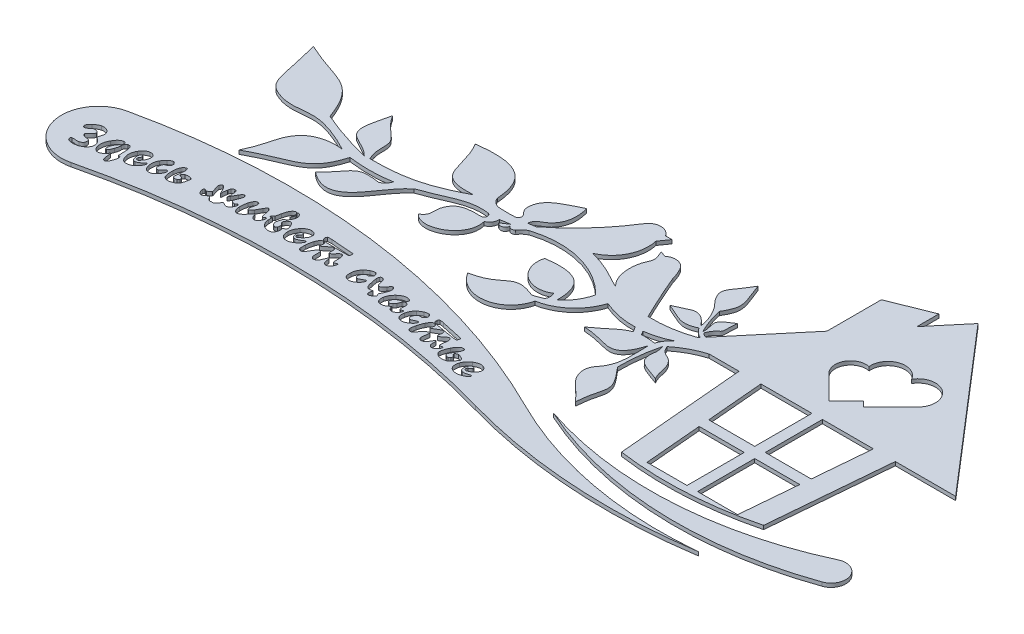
SolidWorks part; units mm, degrees
ref_plane "Спереди" through (0, 0, 0) normal (0, 0, 1) x (1, 0, 0)
ref_plane "Сверху" through (0, 0, 0) normal (0, 1, 0) x (1, 0, 0)
ref_plane "Справа" through (0, 0, 0) normal (1, 0, 0) x (0, 0, -1)
sketch "Эскиз1" plane through (0, 0, 0) normal (0, 1, 0) x (1, 0, 0)
  line L0 (24.9197, 376.2178) -> (1038.9197, 376.2178) construction
  line L1 (-110, -110) -> (110, -110)
  line L2 (-110, -110) -> (-110, 110)
  line L3 (-110, 110) -> (110, 110)
  line L4 (110, -110) -> (110, 110)
  line L5 (-110, -110) -> (110, 110) construction
  line L6 (-110, 110) -> (110, -110) construction
  point P0 (0, 0)
  dimension "D1" = 220
  dimension "D2" = 220
sketch "Эскиз3" plane through (0, 0, 0) normal (0, 1, 0) x (1, 0, 0)
  line L0 (64.2625, 103.9701) -> (64.2625, 60.9701) construction
  line L1 (28.1812, 60.9701) -> (43.3986, 60.9701)
  line L2 (28.1812, 60.9701) -> (45.8403, 82.0154)
  line L3 (64.2625, 103.9701) -> (101.2787, 60.9701)
  line L4 (64.2235, 110.1465) -> (110, 56.9701)
  line L5 (19.6032, 56.9701) -> (39.7333, 56.9701)
  line L6 (19.6032, 56.9701) -> (41.8403, 83.4712)
  line L7 (64.2625, 60.9701) -> (64.2625, 20.5584) construction
  line L8 (62.7625, 60.9701) -> (62.7625, 45.9701)
  line L9 (65.7625, 60.9701) -> (65.7625, 45.9701)
  line L10 (50.7338, 45.9701) -> (62.7625, 45.9701)
  line L11 (50.9963, 42.9701) -> (62.7625, 42.9701)
  line L12 (79.1035, 60.9701) -> (77.7912, 45.9701)
  line L13 (85.1264, 60.9701) -> (82.1276, 26.6936)
  line L14 (52.3086, 27.9701) -> (62.7625, 27.9701)
  line L16 (43.3986, 60.9701) -> (46.5703, 24.7173)
  line L18 (88.7918, 56.9701) -> (86.4291, 29.9651)
  line L19 (19.6032, 56.9701) -> (110, 56.9701) construction
  line L20 (88.7918, 56.9701) -> (110, 56.9701)
  line L21 (62.7625, 60.9701) -> (62.7625, 20.5584) construction
  line L22 (65.7625, 27.9701) -> (76.2164, 27.9701)
  line L23 (65.7625, 60.9701) -> (65.7625, 20.5584) construction
  line L26 (49.4215, 60.9701) -> (62.7625, 60.9701)
  line L27 (28.1812, 60.9701) -> (101.2787, 60.9701) construction
  line L28 (65.7625, 60.9701) -> (79.1035, 60.9701)
  line L29 (85.1264, 60.9701) -> (101.2787, 60.9701)
  line L30 (65.7625, 45.9701) -> (77.7912, 45.9701)
  line L31 (62.7625, 42.9701) -> (62.7625, 27.9701)
  line L32 (65.7625, 42.9701) -> (65.7625, 27.9701)
  line L33 (65.7625, 42.9701) -> (77.5287, 42.9701)
  line L34 (77.5287, 42.9701) -> (76.2164, 27.9701)
  line L35 (39.7333, 56.9701) -> (42.4993, 25.3542)
  line L36 (89.1112, 60.6215) -> (85.1719, 15.5954) construction
  line L37 (39.4138, 60.6215) -> (43.3531, 15.5954) construction
  line L38 (43.3986, 60.9701) -> (85.1264, 60.9701) construction
  line L39 (110, -110) -> (110, 110) construction
  line L40 (45.8403, 82.0154) -> (45.8403, 96.5106)
  line L41 (45.8403, 96.5106) -> (56.9524, 100.9853)
  line L42 (56.9524, 100.9853) -> (56.9524, 95.2583)
  line L43 (56.9524, 95.2583) -> (64.2625, 103.9701)
  line L44 (28.1812, 60.9701) -> (64.2625, 103.9701) construction
  line L45 (41.8403, 83.4712) -> (41.8403, 99.212)
  line L46 (41.8403, 99.212) -> (61.7889, 107.245)
  line L48 (41.8403, 82.0154) -> (41.8403, 99.212) construction
  line L49 (61.7889, 107.245) -> (64.2235, 110.1465)
  line L50 (19.6032, 56.9701) -> (64.2235, 110.1465) construction
  line L51 (41.8403, 99.212) -> (60.9524, 106.9082) construction
  line L52 (60.9524, 106.9082) -> (60.9524, 95.2583) construction
  line L53 (68.2625, 77.8382) -> (68.2625, 69.5358) construction
  line L54 (68.2625, 69.5358) -> (75.4445, 76.7177)
  line L55 (64.2625, 79.8997) -> (72.2625, 79.8997) construction
  line L56 (68.2625, 69.5358) -> (66.9162, 70.8821)
  line L57 (58.805, 75.4277) -> (62.305, 75.4277) construction
  line L58 (62.305, 75.4277) -> (62.305, 66.2709) construction
  line L59 (62.305, 66.2709) -> (55.9766, 72.5993)
  line L60 (62.305, 66.2709) -> (66.9162, 70.8821)
  line L61 (50.9963, 42.9701) -> (52.3086, 27.9701)
  line L62 (49.4215, 60.9701) -> (50.7338, 45.9701)
  line L63 (-110, 7.8444) -> (110, 7.8444) construction
  line L64 (85.1264, 60.9701) -> (81.5066, 19.5954) construction
  line L65 (81.5066, 19.5954) -> (47.0184, 19.5954) construction
  line L66 (43.3986, 60.9701) -> (47.0184, 19.5954) construction
  line L67 (-110, -110) -> (-110, 110) construction
  line L68 (85.1719, 15.5954) -> (43.3531, 15.5954) construction
  line L69 (-99.8714, 39.0204) -> (-91.3859, 20.9097) construction
  arc A0 (68.2625, 81.9613) -> (59.8025, 79.3014) centre (64.2625, 79.8997) ccw
  arc A1 (75.4445, 76.7177) -> (68.2625, 81.9613) centre (72.2625, 79.8997) ccw
  arc A2 (59.8025, 79.3014) -> (55.9766, 72.5993) centre (58.805, 75.4277) ccw
  arc A3 (103.0783, 23.5305) -> (100.051, 30.9259) centre (101.74, 27.3) ccw
  arc A5 (26.6865, 27.4925) -> (100.051, 30.9259) centre (59.1823, 118.6654) ccw
  arc A6 (26.6865, 27.4925) -> (103.0783, 23.5305) centre (69.6614, 117.6558) ccw
  arc A7 (23.1374, 24.7751) -> (83.617, 14.7163) centre (69.6614, 117.6558) ccw
  arc A8 (104.4165, 19.761) -> (98.3621, 34.5519) centre (101.74, 27.3) ccw
  arc A9 (86.4291, 29.9651) -> (98.3621, 34.5519) centre (59.1823, 118.6654) ccw
  arc A10 (28.0294, 31.2604) -> (98.3621, 34.5519) centre (59.1823, 118.6654) ccw construction
  arc A11 (46.5703, 24.7173) -> (82.1276, 26.6936) centre (59.1823, 118.6654) ccw
  arc A12 (27.358, 29.3764) -> (99.2066, 32.7389) centre (59.1823, 118.6654) ccw construction
  arc A13 (24.9654, 23.8817) -> (104.4165, 19.761) centre (69.6614, 117.6558) ccw construction
  arc A14 (23.1374, 24.7751) -> (-97.7946, 39.7277) centre (-58.3735, -137.9539) ccw
  arc A15 (83.617, 14.7163) -> (16.2895, 18.0521) centre (57.1618, 161.8764) cw
  arc A16 (16.2895, 18.0521) -> (-93.282, 20.2443) centre (-42.669, -189.4148) ccw
  arc A17 (-97.7946, 39.7277) -> (-93.282, 20.2443) centre (-95.6286, 29.9651) ccw
  arc A19 (24.9288, 28.3515) -> (-98.661, 43.6327) centre (-58.3735, -137.9539) ccw
  arc A20 (-98.661, 43.6327) -> (-92.3433, 16.356) centre (-95.6286, 29.9651) ccw
  arc A21 (15.1961, 14.2044) -> (-92.3433, 16.356) centre (-42.669, -189.4148) ccw
  point P4 (64.2625, 60.9701)
  dimension "D12" = 9
  dimension "D15" = 8
  dimension "D20" = 8
  dimension "D23" = 20
  dimension "D1" = 40
  dimension "D2" = 43
  dimension "D6" = 3
  dimension "D7" = 5
  dimension "D8" = 15
  dimension "D9" = 15
  dimension "D13" = 8
  dimension "D14" = 45
  dimension "D16" = 3.5
  dimension "D17" = 45
  dimension "D18" = 6
  dimension "D3" = 4
  dimension "D4" = 1.5
  dimension "D5" = 1.5
  dimension "D10" = 4
  dimension "D11" = 4
  dimension "D19" = 4
  dimension "D21" = 4
  dimension "D22" = 2
  dimension "D24" = 4
sketch "Эскиз4" plane through (0, 0, 0) normal (0, 1, 0) x (1, 0, 0)
  line L0 (-70, 8.9797) -> (70, 8.9797) construction
  line L1 (-66.276, 48.806) -> (66.4656, 48.8233)
  line L3 (0, 0) -> (0, 8.9797) construction
  arc A0 (-66.276, 48.806) -> (-61.7647, -30.1633) centre (-70, 8.9797) ccw
  arc A1 (-98.9066, 22.9467) -> (18.8733, 19.0244) centre (-47.3155, -198.186) cw construction
  arc A2 (17.3829, 21.8997) -> (-94.2206, 24.1326) centre (-42.669, -189.4148) ccw
  arc A3 (20.3824, 21.0242) -> (-98.9066, 22.9467) centre (-42.669, -189.4148) ccw construction
  arc A4 (61.7647, -30.1633) -> (66.4656, 48.8233) centre (70, 8.9797) ccw
  arc A5 (-61.7647, -30.1633) -> (61.7647, -30.1633) centre (0, -323.7364) cw
  point P10 (1.414, 12.964)
  dimension "D3" = 40
  dimension "D4" = 40
  dimension "D5" = 300
  dimension "D2" = 140
  dimension "D1" = 4
sketch "Эскиз5" plane through (0, 0, 0) normal (0, 1, 0) x (1, 0, 0)
  line L0 (19.4678, 57.3611) -> (20.1869, 56.1334)
  line L1 (21.4931, 57.5238) -> (22.1246, 56.5168)
  line L2 (7.1547, 77.7869) -> (5.5048, 78.3997)
  line L3 (5.5048, 78.3997) -> (6.2156, 76.5198)
  line L4 (2.6024, 79.9565) -> (4.4345, 82.5645)
  line L5 (4.4345, 82.5645) -> (2.6024, 82.5645)
  line L6 (32.6801, 75.9406) -> (38.6301, 79.2463)
  line L7 (-77.7166, 47.1129) -> (-78.2226, 46.1222)
  arc A0 (27.6672, 56.3188) -> (26.4504, 45.966) centre (67.0603, 46.4409) ccw
  arc A1 (28.3849, 57.1795) -> (38.4245, 61.6181) centre (41.6095, 40.8401) cw
  arc A2 (25.8064, 56.3188) -> (29.1303, 60.128) centre (31.504, 54.7019) cw
  arc A3 (29.1303, 60.128) -> (21.4931, 57.5238) centre (18.8463, 77.7869) cw
  arc A4 (19.4678, 57.3611) -> (10.5596, 59.1073) centre (18.8463, 77.7869) cw
  arc A5 (4.8332, 65.6803) -> (7.1547, 64.4869) centre (19.9633, 92.2585) ccw
  arc A6 (30.5687, 63.5732) -> (28.1974, 65.5826) centre (32.4248, 68.1674) cw
  arc A7 (30.1155, 65.2643) -> (31.2408, 64.6261) centre (31.5857, 66.5456) ccw
  arc A8 (27.1889, 72.2037) -> (29.4866, 65.6803) centre (55.1893, 78.3997) ccw
  arc A9 (27.822, 66.762) -> (25.2436, 72.6741) centre (14.8033, 64.6025) ccw
  arc A10 (18.8463, 61.6959) -> (13.422, 73.6764) centre (232.08, 165.4576) cw
  arc A11 (7.1547, 77.7869) -> (12.1628, 76.8463) centre (9.266, 75.2251) cw
  arc A12 (12.1628, 76.8463) -> (13.422, 73.6764) centre (0.8643, 70.5231) cw
  arc A13 (18.8463, 61.6959) -> (30.5687, 63.5732) centre (19.9633, 92.2585) ccw
  arc A14 (4.8332, 65.6803) -> (-2.8095, 68.8088) centre (-11.0495, 37.7801) ccw
  arc A15 (-16.7249, 65.4567) -> (6.7404, 59.5803) centre (-9.7268, 43.6133) cw
  arc A16 (-2.8095, 68.8088) -> (2.6024, 79.9565) centre (-7.0292, 77.7449) ccw
  arc A17 (2.6024, 82.5645) -> (-3.1371, 82.5593) centre (-0.2657, 80.7486) ccw
  arc A18 (-3.1371, 82.5593) -> (-16.794, 67.4541) centre (-53.321, 114.2051) cw
  arc A19 (-22.757, 63.3551) -> (-20.2996, 63.7937) centre (-21.6147, 64.0583) ccw
  arc A20 (-20.2996, 63.7937) -> (-18.6001, 63.7937) centre (-19.4499, 64.6435) ccw
  arc A21 (-16.7249, 65.4567) -> (-18.6001, 63.7937) centre (-14.7474, 61.3381) ccw
  arc A22 (-23.1659, 64.0583) -> (-21.0561, 64.417) centre (-15.623, 26.0783) cw
  arc A23 (-25.7505, 66.9301) -> (-21.8358, 66.9301) centre (-23.7932, 110.2778) ccw
  arc A24 (-21.0561, 64.417) -> (-22.757, 63.3551) centre (-53.321, 114.2051) cw
  arc A25 (0.2898, 50.01) -> (10.5596, 59.1073) centre (-2.3445, 63.3292) ccw
  arc A26 (6.7404, 59.5803) -> (2.9913, 53.4771) centre (-4.13, 62.0547) cw
  arc A27 (6.9888, 82.1815) -> (15.6533, 78.7998) centre (9.266, 75.2251) cw
  arc A28 (15.6533, 78.7998) -> (17.2194, 74.9649) centre (0.8643, 70.5231) cw
  arc A29 (18.7732, 71.3609) -> (17.2194, 74.9649) centre (232.08, 165.4576) cw
  arc A30 (22.4431, 63.4461) -> (17.2194, 74.9649) centre (232.08, 165.4576) cw construction
  arc A31 (-18.6001, 67.1978) -> (-16.794, 67.4541) centre (-23.7932, 110.2778) ccw
  arc A32 (6.9888, 82.1815) -> (-6.5206, 84.6929) centre (-0.2657, 80.7486) ccw
  arc A33 (-6.5206, 84.6929) -> (-10.2784, 79.4404) centre (-53.321, 114.2051) cw
  arc A34 (-6.5206, 84.6929) -> (-19.2567, 70.6061) centre (-53.321, 114.2051) cw construction
  arc A35 (5.982, 84.7042) -> (-6.5206, 84.6929) centre (-0.2657, 80.7486) ccw construction
  arc A36 (4.6108, 80.8737) -> (15.6533, 78.7998) centre (9.266, 75.2251) cw construction
  arc A37 (-15.327, 47.7127) -> (0.2898, 50.01) centre (-7.9678, 51.9148) ccw
  arc A38 (-8.3753, 61.3381) -> (0.8643, 54.2489) centre (-2.4156, 59.5399) ccw
  arc A39 (0.8643, 54.2489) -> (0.8643, 52.0875) centre (-1.2063, 53.1682) cw
  arc A40 (0.8643, 52.0875) -> (-1.6675, 51.1816) centre (-4.13, 62.0547) cw
  arc A41 (-25.7505, 66.9301) -> (-28.3732, 68.8088) centre (-25.6673, 69.8162) cw
  arc A42 (-26.3597, 64.0583) -> (-26.581, 62.5386) centre (-26.4704, 63.2985) cw
  arc A43 (-23.1659, 64.0583) -> (-24.7346, 61.6181) centre (-25.7573, 63.9998) cw
  arc A44 (-47.9015, 56.7778) -> (-46.1807, 58.622) centre (-49.077, 59.5994) ccw
  arc A45 (-56.2461, 61.045) -> (-69.4638, 65.4567) centre (-37.2613, 139.9298) cw
  spline S0 degree 3 poles (28.864, 31.9915) (29.1088, 36.1758) (30.1262, 38.2083) (30.1196, 41.0626) (29.3386, 42.6134) (26.4504, 45.966) knots 0 0 0 0 0.448203 0.548203 1 1 1 1
  spline S1 degree 3 poles (25.4671, 54.2489) (25.5173, 50.6569) (25.6797, 49.6888) (25.1124, 46.3323) (24.3246, 44.441) (22.0407, 41.7038) (22.9149, 36.5797) (26.4478, 35.1323) (28.864, 31.9915) knots 0 0 0 0 0.262515 0.304969 0.411252 0.445475 0.633918 1 1 1 1
  spline S2 degree 3 poles (27.6672, 56.3188) (28.3045, 53.9957) (27.2385, 53.4399) (28.6078, 50.1196) (30.5333, 49.3866) (34.3409, 48.063) knots 0 0 0 0 0.587102 0.687102 1 1 1 1
  spline S3 degree 3 poles (28.3849, 57.1795) (29.1923, 54.9931) (30.8853, 55.4261) (33.5762, 51.8287) (32.9236, 50.2449) (34.3409, 48.063) knots 0 0 0 0 0.398325 0.498325 1 1 1 1
  spline S4 degree 2 poles (25.4671, 54.2489) (25.6465, 53.3545) (25.4982, 52.6234) knots 0 0 0 0.045717 0.045717 0.045717
  spline S5 degree 3 poles (12.4577, 50.651) (17.1173, 50.4382) (20.581, 48.0281) (24.2467, 50.5319) (25.4671, 54.2489) knots 0 0 0 0 0.57212 1 1 1 1
  spline S6 degree 2 poles (25.8064, 56.3188) (23.6043, 56.6296) (22.1246, 56.5168) knots 0 0 0 0.2017 0.2017 0.2017
  spline S7 degree 3 poles (20.1869, 56.1334) (19.9461, 56.0505) (19.4858, 55.8613) (17.3232, 54.6994) (15.6338, 52.8537) (12.4577, 50.651) knots 0.353395 0.353395 0.353395 0.353395 0.417809 0.482469 1 1 1 1
  spline S8 degree 3 poles (30.1155, 65.2643) (30.7673, 67.1396) (32.8462, 67.7574) (32.0339, 69.5856) (32.4248, 72.0657) knots 0 0 0 0 0.440299 1 1 1 1
  spline S9 degree 3 poles (29.4866, 65.6803) (29.5495, 66.918) (28.7194, 68.5444) (29.6678, 70.4068) (30.3583, 70.6308) (32.4248, 72.0657) knots 0 0 0 0 0.392131 0.492131 1 1 1 1
  spline S10 degree 3 poles (27.1889, 72.2037) (28.6875, 74.7307) (28.9636, 77.5082) (27.6486, 80.2711) (26.4504, 83.4163) knots 0 0 0 0 0.437978 1 1 1 1
  spline S11 degree 3 poles (26.4504, 83.4163) (24.5288, 79.9961) (21.0811, 77.0285) (24.2801, 73.6675) (25.2436, 72.6741) knots 0 0 0 0 0.439909 1 1 1 1
  spline S12 degree 3 poles (27.822, 66.762) (26.36, 68.5846) (23.5856, 69.9175) (21.8685, 68.2115) (18.8463, 67.0583) knots 0 0 0 0 0.435142 1 1 1 1
  spline S13 degree 3 poles (28.1974, 65.5826) (24.1965, 63.8319) (23.3678, 65.3547) (18.8463, 67.0583) knots 0 0 0 0 1 1 1 1
  spline S14 degree 3 poles (6.2156, 76.5198) (6.613, 75.2328) (4.5903, 72.3616) (4.9375, 66.7491) (7.1547, 64.4869) knots 0 0 0 0 0.212545 1 1 1 1
  spline S15 degree 1 poles (30.6294, 70.1633) (27.1473, 92.823) knots 0 0 1 1 construction
  spline S16 degree 1 poles (27.1473, 92.823) (22.3722, 69.8893) knots 0 0 1 1 construction
  spline S17 degree 3 poles (30.6294, 70.1633) (30.8052, 70.4597) (31.1548, 71.075) (31.7297, 72.2071) (32.2875, 73.5781) (32.6706, 75.2341) (32.7108, 76.5624) (32.6251, 77.4728) (32.505, 78.2509) (32.1997, 79.5706) (31.5924, 81.2775) (30.8431, 83.1384) (30.1036, 85.0597) (29.3057, 87.1591) (28.3284, 89.7219) (27.5405, 91.7909) (27.1473, 92.823) knots 0 0 0 0 0.046109 0.092218 0.184435 0.276653 0.36887 0.414979 0.461088 0.553306 0.737741 0.922176 1.014394 1.106611 1.291046 1.475482 1.475482 1.475482 1.475482 only from (32.6801, 75.9406) to (27.1473, 92.823)
  spline S18 degree 3 poles (27.1473, 92.823) (26.7871, 92.1819) (26.0669, 90.9) (24.9858, 88.9758) (24.0869, 87.376) (23.4538, 86.2489) (23.1425, 85.6952) (22.9562, 85.363) (22.7285, 84.9613) (22.3766, 84.37) (21.7954, 83.456) (21.1153, 82.4708) (20.3532, 81.3997) (19.7074, 80.4026) (19.2117, 79.3629) (18.8991, 78.4226) (18.7333, 77.3369) (18.7597, 75.9937) (19.1132, 74.5438) (19.7571, 73.1771) (20.4753, 72.0694) (21.1967, 71.1574) (21.748, 70.5432) (22.1379, 70.1313) (22.2903, 69.9737) (22.3722, 69.8893) knots -0.319292 -0.319292 -0.319292 -0.319292 -0.236836 -0.154381 -0.071925 -0.030697 -0.010083 0.000224 0.010531 0.051759 0.092987 0.175442 0.257898 0.340354 0.381582 0.42281 0.464038 0.505265 0.587721 0.670177 0.752633 0.835088 0.917544 0.958772 1 1 1 1 only from (27.1473, 92.823) to (20.4307, 72.1657)
  spline S19 degree 1 poles (30.9423, 69.2647) (17.4203, 70.7955) knots 0 0 1 1 construction
  spline S20 degree 3 poles (30.9423, 69.2647) (30.6812, 69.5902) (30.1248, 70.2352) (28.9969, 71.3332) (27.4391, 72.4464) (25.2385, 73.2112) (23.3591, 73.186) (22.0829, 72.8677) (21.042, 72.475) (20.2646, 72.0842) (19.512, 71.7093) (18.9122, 71.421) (18.3457, 71.1684) (17.8415, 70.9594) (17.5587, 70.8483) (17.4203, 70.7955) knots 0 0 0 0 0.0625 0.125 0.25 0.375 0.5 0.5625 0.625 0.75 0.8125 0.875 0.9375 0.96875 1 1 1 1 only from (20.4307, 72.1657) to (18.7732, 71.3609)
  spline S21 degree 3 poles (-18.6001, 67.1978) (-18.2274, 69.3391) (-15.8629, 68.7074) (-13.2684, 74.0361) (-13.6602, 76.7101) (-14.141, 78.3997) knots 0 0 0 0 0.560438 0.660438 1 1 1 1
  spline S22 degree 3 poles (-14.141, 78.3997) (-17.4129, 76.7273) (-21.8781, 75.2141) (-22.7538, 69.3543) (-20.55, 68.3378) (-21.1817, 67.0782) (-21.8358, 66.9301) knots 0 0 0 0 0.452436 0.534421 0.788133 1 1 1 1
  spline S23 degree 1 poles (-14.8622, 65.7737) (-11.6263, 84.1774) knots 0 0 1 1 construction
  spline S24 degree 1 poles (-11.6263, 84.1774) (-25.7505, 67.7514) knots 0 0 1 1 construction
  spline S25 degree 3 poles (-14.8622, 65.7737) (-14.7576, 65.8356) (-14.567, 65.9489) (-14.0459, 66.2751) (-13.2758, 66.8236) (-12.2735, 67.7642) (-11.3374, 68.9898) (-10.5598, 70.4077) (-9.9439, 72.1081) (-9.6531, 73.7974) (-9.6017, 75.3881) (-9.7229, 76.8692) (-9.9242, 78.0115) (-10.1169, 78.8475) (-10.2891, 79.4845) (-10.4169, 79.9254) (-10.598, 80.5645) (-10.8207, 81.3458) (-11.179, 82.6057) (-11.4473, 83.5484) (-11.6263, 84.1774) knots 0.302463 0.302463 0.302463 0.302463 0.334065 0.365666 0.428869 0.492072 0.555275 0.618478 0.681681 0.744884 0.808086 0.871289 0.934492 0.966094 0.997695 1.029297 1.060898 1.124101 1.187304 1.31371 1.31371 1.31371 1.31371 only from (-10.2784, 79.4404) to (-11.6263, 84.1774)
  spline S26 degree 3 poles (-11.6263, 84.1774) (-12.3638, 83.8004) (-13.4737, 83.2326) (-14.9387, 82.4851) (-15.8852, 81.9977) (-16.5426, 81.6696) (-17.2635, 81.3209) (-18.5921, 80.69) (-20.6525, 79.6665) (-22.7856, 78.261) (-24.3903, 76.6407) (-25.4392, 75.1292) (-26.1879, 73.2584) (-26.4487, 71.7488) (-26.4743, 70.4534) (-26.3586, 69.4701) (-26.1074, 68.5418) (-25.8827, 68.0142) (-25.7505, 67.7514) knots -0.199828 -0.199828 -0.199828 -0.199828 -0.097852 -0.046863 0.004125 0.029619 0.055113 0.106101 0.208077 0.310053 0.361041 0.412029 0.463017 0.514005 0.539499 0.564993 0.590487 0.615981 0.615981 0.615981 0.615981 only from (-11.6263, 84.1774) to (-25.5338, 74.788)
  spline S27 degree 3 poles (-15.327, 47.7127) (-7.0902, 49.258) (-9.1779, 54.2284) (-1.6675, 51.1816) knots 0 0 0 0 1 1 1 1
  spline S28 degree 3 poles (2.9913, 53.4771) (2.9279, 59.9836) (0.1931, 62.5241) (-8.3753, 61.3381) knots 0 0 0 0 1 1 1 1
  spline S29 degree 3 poles (-44.0346, 78.3997) (-31.4187, 80.2501) (-28.9075, 75.4359) (-28.3732, 68.8088) knots 0 0 0 0 1 1 1 1
  spline S30 degree 3 poles (-44.0346, 78.3997) (-39.6734, 71.372) (-43.0205, 65.6475) (-32.8408, 66.2981) knots 0 0 0 0 1 1 1 1
  spline S31 degree 3 poles (-32.8408, 66.2981) (-40.4611, 62.364) (-45.409, 60.972) (-54.4339, 61.045) knots 0 0 0 0 1 1 1 1
  spline S32 degree 3 poles (-57.3626, 58.4909) (-52.8684, 57.9059) (-49.2421, 58.0726) (-46.1807, 58.622) knots 0 0 0 0 0.256014 0.256014 0.256014 0.256014
  spline S33 degree 1 poles (-43.3924, 66.2308) (-54.4016, 65.0449) knots 0 0 1 1 construction
  spline S34 degree 1 poles (-50.6491, 81.4724) (-43.3924, 66.2308) knots 0 0 1 1 construction
  spline S35 degree 1 poles (-50.6491, 81.4724) (-24.3861, 69.1303) knots 0 0 1 1 construction
  spline S36 degree 3 poles (-54.4016, 65.0449) (-53.8419, 65.0403) (-52.6941, 65.0435) (-50.6251, 65.1026) (-48.2695, 65.2759) (-45.7476, 65.649) (-44.1784, 66.0135) (-43.3924, 66.2308) knots 0.460482 0.460482 0.460482 0.460482 0.527922 0.595362 0.730241 0.865121 1 1 1 1 only from (-51.3001, 65.0886) to (-43.3924, 66.2308)
  spline S37 degree 3 poles (-43.3924, 66.2308) (-43.6194, 66.567) (-44.0387, 67.2933) (-44.6298, 68.6455) (-45.1235, 70.2283) (-45.5964, 71.9677) (-46.0317, 73.3498) (-46.4623, 74.4393) (-46.7799, 75.1234) (-47.0671, 75.6691) (-47.2716, 76.0264) (-47.4285, 76.2834) (-47.6705, 76.6722) (-48.0543, 77.2913) (-48.6232, 78.2078) (-49.5219, 79.6561) (-50.1986, 80.7464) (-50.6491, 81.4724) knots -0.245781 -0.245781 -0.245781 -0.245781 -0.19413 -0.14248 -0.039179 0.064122 0.167422 0.219073 0.270723 0.296548 0.322373 0.335286 0.348199 0.374024 0.425674 0.477324 0.580625 0.580625 0.580625 0.580625
  spline S38 degree 3 poles (-50.6491, 81.4724) (-49.7349, 81.6064) (-48.3637, 81.8074) (-46.5349, 82.076) (-45.3932, 82.2425) (-44.4769, 82.3789) (-43.4816, 82.5151) (-41.8444, 82.6981) (-39.6351, 82.83) (-37.2097, 82.7702) (-34.2241, 82.3895) (-30.8973, 81.2994) (-27.7096, 78.8487) (-25.7303, 75.6812) (-24.7468, 72.3852) (-24.4744, 70.2254) (-24.3861, 69.1303) knots -0.159428 -0.159428 -0.159428 -0.159428 -0.086964 -0.050731 -0.014499 0.003617 0.021733 0.057965 0.130429 0.202893 0.275358 0.420286 0.565215 0.710143 0.855072 1 1 1 1 only from (-50.6491, 81.4724) to (-25.5338, 74.788)
  spline S39 degree 3 poles (-35.4507, 54.7019) (-32.458, 50.8459) (-23.2533, 55.0728) (-24.7346, 61.6181) knots 0 0 0 0 1 1 1 1
  spline S40 degree 3 poles (-26.581, 62.5386) (-29.4845, 62.616) (-32.196, 62.3195) (-34.8092, 57.5268) (-33.1149, 56.1296) (-35.4507, 54.7019) knots 0 0 0 0 0.380693 0.480693 1 1 1 1
  spline S41 degree 3 poles (-58.8182, 50.651) (-55.9302, 53.2618) (-54.3551, 57.1374) (-50.7365, 57.1618) (-47.9015, 56.7778) knots 0 0 0 0 0.597042 1 1 1 1
  spline S42 degree 3 poles (-58.8182, 50.651) (-52.8866, 45.927) (-47.8378, 51.4987) (-43.6472, 58.0811) (-41.6311, 59.8012) knots 0 0 0 0 0.68526 1 1 1 1
  spline S43 degree 3 poles (-41.6311, 59.8012) (-35.6429, 61.825) (-31.8828, 64.8627) (-26.3597, 64.0583) knots 0.395484 0.395484 0.395484 0.395484 1 1 1 1
  spline S44 degree 3 poles (-61.4061, 74.1485) (-59.3121, 70.3906) (-53.9826, 68.5912) (-55.7567, 63.7995) (-54.4339, 61.045) knots 0 0 0 0 0.593908 1 1 1 1
  spline S45 degree 3 poles (-61.4061, 74.1485) (-62.4592, 69.6187) (-64.3272, 64.1557) (-58.1897, 62.8667) (-56.2461, 61.045) knots 0 0 0 0 0.586984 1 1 1 1
  spline S46 degree 3 poles (-69.4638, 65.4567) (-73.7379, 76.9363) (-77.325, 74.388) (-87.9656, 79.4404) knots 0 0 0 0 1 1 1 1
  spline S47 degree 3 poles (-87.9656, 79.4404) (-85.4912, 69.9878) (-85.8568, 65.5282) (-77.3942, 61.8858) (-71.6532, 64.8855) (-63.0226, 60.755) (-60.8673, 59.5994) knots 0 0 0 0 0.258742 0.329402 0.664695 1 1 1 1
  spline S48 degree 3 poles (-57.3626, 58.4909) (-60.0804, 49.2999) (-64.4518, 50.7723) (-74.1544, 45.2932) knots 0 0 0 0 1 1 1 1
  spline S49 degree 3 poles (-60.8673, 59.5994) (-66.849, 60.0678) (-71.9927, 54.9872) (-71.8443, 49.8157) (-74.1544, 45.2932) knots 0 0 0 0 0.525603 1 1 1 1
  spline S50 degree 1 poles (-62.9558, 85.1473) (-58.9815, 58.1265) knots 0 0 1 1 construction
  spline S51 degree 1 poles (-62.9558, 85.1473) (-50.8281, 62.7766) knots 0 0 1 1 construction
  spline S52 degree 3 poles (-58.9815, 58.1265) (-59.0911, 58.2293) (-59.312, 58.4148) (-59.867, 58.8032) (-60.7444, 59.29) (-61.8545, 59.8284) (-62.8795, 60.3874) (-63.719, 60.9246) (-64.6315, 61.6682) (-65.797, 63.0425) (-66.6141, 65.0109) (-66.8088, 67.1804) (-66.635, 69.1115) (-66.2835, 70.9604) (-65.8387, 72.8301) (-65.3708, 74.7404) (-64.727, 77.5393) (-63.9218, 80.988) (-63.2778, 83.7622) (-62.9558, 85.1473) knots -0.435964 -0.435964 -0.435964 -0.435964 -0.39109 -0.346216 -0.256469 -0.166721 -0.121847 -0.076973 -0.032099 0.012775 0.102522 0.19227 0.282018 0.371766 0.461513 0.551261 0.641009 0.820504 1 1 1 1 only from (-66.6073, 69.0836) to (-62.9558, 85.1473)
  spline S53 degree 3 poles (-62.9558, 85.1473) (-62.3049, 83.9792) (-61.3286, 82.2271) (-60.1895, 80.1829) (-59.5387, 79.0149) (-59.0504, 78.1386) (-58.644, 77.4092) (-58.3178, 76.8238) (-58.1163, 76.4622) (-57.9704, 76.2005) (-57.8947, 76.0644) (-57.8186, 75.9307) (-57.6278, 75.6132) (-57.218, 75.0186) (-56.5628, 74.2548) (-55.6633, 73.4044) (-54.6326, 72.5131) (-53.6562, 71.6149) (-52.8309, 70.6503) (-52.23, 69.7572) (-51.71, 68.6439) (-51.4135, 67.4205) (-51.327, 66.4665) (-51.3011, 65.4384) (-51.2987, 64.5334) (-51.2072, 63.8501) (-51.0514, 63.2915) (-50.9057, 62.9381) (-50.8281, 62.7766) knots -0.476854 -0.476854 -0.476854 -0.476854 -0.292247 -0.199944 -0.153792 -0.107641 -0.061489 -0.038413 -0.015337 -0.003799 0.00197 0.007739 0.030814 0.076966 0.16927 0.261573 0.353876 0.44618 0.492331 0.538483 0.584635 0.630786 0.676938 0.72309 0.815393 0.907697 0.953848 1 1 1 1 only from (-62.9558, 85.1473) to (-51.3001, 65.0886)
  spline S54 degree 1 poles (-65.7151, 66.8525) (-94.0108, 86.7388) knots 0 0 1 1 construction
  spline S55 degree 1 poles (-94.0108, 86.7388) (-72.6438, 59.2183) knots 0 0 1 1 construction
  spline S56 degree 1 poles (-72.6438, 59.2183) (-77.7166, 47.1129) knots 0 0 1 1 construction
  spline S57 degree 3 poles (-65.7151, 66.8525) (-65.888, 67.3166) (-66.2544, 68.2614) (-66.9771, 69.9591) (-67.922, 71.8691) (-69.1593, 73.8447) (-70.5517, 75.5439) (-72.1038, 76.952) (-74.3124, 78.4243) (-77.0975, 79.5983) (-79.8706, 80.5025) (-82.3117, 81.3732) (-83.9691, 82.0288) (-85.229, 82.58) (-85.9661, 82.9185) (-86.7679, 83.3) (-87.8134, 83.796) (-90.2869, 84.9707) (-92.3574, 85.9537) (-94.0108, 86.7388) knots 0 0 0 0 0.038848 0.077695 0.15539 0.233086 0.310781 0.388476 0.466171 0.621562 0.776952 0.854647 0.932342 0.97119 0.990614 1.010038 1.048885 1.087733 1.243123 1.243123 1.243123 1.243123 only from (-66.6073, 69.0836) to (-94.0108, 86.7388)
  spline S58 degree 3 poles (-94.0108, 86.7388) (-93.6098, 85.2068) (-93.0071, 82.9048) (-92.3081, 80.2331) (-91.9027, 78.6866) (-91.3279, 76.4774) (-90.6672, 73.6179) (-90.0233, 70.5129) (-89.4695, 67.9406) (-88.8123, 65.6271) (-87.8561, 63.6753) (-86.6667, 62.2456) (-85.2235, 61.0223) (-83.3674, 60.0747) (-81.377, 59.4024) (-79.489, 59.0114) (-77.1519, 58.8241) (-75.1883, 58.9777) (-73.8235, 59.1244) (-73.1219, 59.188) (-72.8063, 59.2098) (-72.6438, 59.2183) knots -0.075834 -0.075834 -0.075834 -0.075834 -0.0339 -0.012933 -0.002449 0.008035 0.049969 0.091904 0.133838 0.175772 0.217707 0.238674 0.259641 0.301576 0.34351 0.385445 0.427379 0.511248 0.553183 0.57415 0.595117 0.595117 0.595117 0.595117
  spline S59 degree 3 poles (-72.6438, 59.2183) (-72.8636, 58.955) (-73.2864, 58.4001) (-73.9918, 57.2965) (-74.6697, 55.9103) (-75.2063, 54.3579) (-75.5842, 52.9665) (-75.9235, 51.6743) (-76.3184, 50.3631) (-76.7755, 49.1365) (-77.2572, 48.041) (-77.5634, 47.4128) (-77.7166, 47.1129) knots 0.395215 0.395215 0.395215 0.395215 0.433014 0.470813 0.546412 0.62201 0.697608 0.773206 0.848804 0.924402 0.962201 1 1 1 1
  dimension "D1" = 4
  dimension "D2" = 4
  dimension "D3" = 4
  dimension "D4" = 4
  dimension "D5" = 4
  dimension "D6" = 4
  dimension "D7" = 4
  dimension "D8" = 4
sketch "Эскиз13" plane through (0, 0, 0) normal (0, 1, 0) x (1, 0, 0)
  line L65 (82.1276, 26.6936) -> (85.1264, 60.9701)
  line L66 (85.1264, 60.9701) -> (101.2787, 60.9701)
  line L67 (101.2787, 60.9701) -> (64.2625, 103.9701)
  line L68 (64.2625, 103.9701) -> (56.9524, 95.2583)
  line L69 (56.9524, 95.2583) -> (56.9524, 100.9853)
  line L70 (56.9524, 100.9853) -> (45.8403, 96.5106)
  line L71 (45.8403, 96.5106) -> (45.8403, 82.0154)
  line L72 (45.8403, 82.0154) -> (28.1812, 60.9701)
  line L73 (28.1812, 60.9701) -> (43.3986, 60.9701)
  line L74 (43.3986, 60.9701) -> (46.5703, 24.7173)
  line L75 (82.3122, 28.8036) -> (85.1264, 60.9701)
  line L76 (85.1264, 60.9701) -> (101.2787, 60.9701)
  line L77 (101.2787, 60.9701) -> (64.2625, 103.9701)
  line L78 (64.2625, 103.9701) -> (56.9524, 95.2583)
  line L79 (56.9524, 95.2583) -> (56.9524, 100.9853)
  line L80 (56.9524, 100.9853) -> (45.8403, 96.5106)
  line L81 (45.8403, 96.5106) -> (45.8403, 82.0154)
  line L82 (30.4187, 63.6366) -> (30.2761, 63.4667)
  line L83 (35.5555, 60.9701) -> (43.3986, 60.9701)
  line L84 (43.3986, 60.9701) -> (46.3916, 26.7603)
  line L89 (55.9766, 72.5993) -> (62.305, 66.2709)
  line L90 (62.305, 66.2709) -> (66.9162, 70.8821)
  line L91 (66.9162, 70.8821) -> (68.2625, 69.5358)
  line L92 (68.2625, 69.5358) -> (75.4445, 76.7177)
  line L93 (55.9766, 72.5993) -> (62.305, 66.2709)
  line L94 (62.305, 66.2709) -> (66.9162, 70.8821)
  line L95 (66.9162, 70.8821) -> (68.2625, 69.5358)
  line L96 (68.2625, 69.5358) -> (75.4445, 76.7177)
  line L163 (62.7625, 42.9701) -> (50.9963, 42.9701)
  line L164 (62.7625, 27.9701) -> (62.7625, 42.9701)
  line L165 (52.3086, 27.9701) -> (62.7625, 27.9701)
  line L166 (50.9963, 42.9701) -> (52.3086, 27.9701)
  line L167 (62.7625, 42.9701) -> (50.9963, 42.9701)
  line L168 (62.7625, 27.9701) -> (62.7625, 42.9701)
  line L169 (52.3086, 27.9701) -> (62.7625, 27.9701)
  line L170 (50.9963, 42.9701) -> (52.3086, 27.9701)
  line L181 (65.7625, 42.9701) -> (65.7625, 27.9701)
  line L182 (65.7625, 27.9701) -> (76.2164, 27.9701)
  line L183 (76.2164, 27.9701) -> (77.5287, 42.9701)
  line L184 (77.5287, 42.9701) -> (65.7625, 42.9701)
  line L185 (65.7625, 42.9701) -> (65.7625, 27.9701)
  line L186 (65.7625, 27.9701) -> (76.2164, 27.9701)
  line L187 (76.2164, 27.9701) -> (77.5287, 42.9701)
  line L188 (77.5287, 42.9701) -> (65.7625, 42.9701)
  line L199 (65.7625, 45.9701) -> (77.7912, 45.9701)
  line L200 (77.7912, 45.9701) -> (79.1035, 60.9701)
  line L201 (79.1035, 60.9701) -> (65.7625, 60.9701)
  line L202 (65.7625, 60.9701) -> (65.7625, 45.9701)
  line L203 (65.7625, 45.9701) -> (77.7912, 45.9701)
  line L204 (77.7912, 45.9701) -> (79.1035, 60.9701)
  line L205 (79.1035, 60.9701) -> (65.7625, 60.9701)
  line L206 (65.7625, 60.9701) -> (65.7625, 45.9701)
  line L217 (49.4215, 60.9701) -> (50.7338, 45.9701)
  line L218 (50.7338, 45.9701) -> (62.7625, 45.9701)
  line L219 (62.7625, 45.9701) -> (62.7625, 60.9701)
  line L220 (62.7625, 60.9701) -> (49.4215, 60.9701)
  line L221 (49.4215, 60.9701) -> (50.7338, 45.9701)
  line L222 (50.7338, 45.9701) -> (62.7625, 45.9701)
  line L223 (62.7625, 45.9701) -> (62.7625, 60.9701)
  line L224 (62.7625, 60.9701) -> (49.4215, 60.9701)
  line L226 (22.1246, 56.5168) -> (21.4931, 57.5238)
  line L227 (22.1246, 56.5168) -> (21.4931, 57.5238)
  line L249 (20.1869, 56.1334) -> (19.4678, 57.3611)
  line L250 (20.1869, 56.1334) -> (19.4678, 57.3611)
  line L280 (45.8403, 82.0154) -> (31.2479, 64.6248)
  line L284 (7.1547, 77.7869) -> (5.5048, 78.3997)
  line L285 (5.5048, 78.3997) -> (6.2156, 76.5198)
  line L286 (2.6024, 79.9565) -> (4.4345, 82.5645)
  line L287 (4.4345, 82.5645) -> (2.6024, 82.5645)
  line L288 (7.1547, 77.7869) -> (5.5048, 78.3997)
  line L289 (5.5048, 78.3997) -> (6.2156, 76.5198)
  line L290 (2.6024, 79.9565) -> (4.4345, 82.5645)
  line L291 (4.4345, 82.5645) -> (2.6024, 82.5645)
  arc A20 (16.2895, 18.0521) -> (83.617, 14.7163) centre (57.1618, 161.8764) ccw
  arc A21 (23.1374, 24.7751) -> (83.617, 14.7163) centre (69.6614, 117.6558) ccw
  arc A22 (16.2895, 18.0521) -> (-93.282, 20.2443) centre (-42.669, -189.4148) ccw
  arc A23 (-97.7946, 39.7277) -> (-93.282, 20.2443) centre (-95.6286, 29.9651) ccw
  arc A24 (23.1374, 24.7751) -> (-97.7946, 39.7277) centre (-58.3735, -137.9539) ccw
  arc A25 (16.2895, 18.0521) -> (83.617, 14.7163) centre (57.1618, 161.8764) ccw
  arc A26 (23.1374, 24.7751) -> (83.617, 14.7163) centre (69.6614, 117.6558) ccw
  arc A27 (16.2895, 18.0521) -> (-93.282, 20.2443) centre (-42.669, -189.4148) ccw
  arc A28 (-97.7946, 39.7277) -> (-93.282, 20.2443) centre (-95.6286, 29.9651) ccw
  arc A29 (23.1374, 24.7751) -> (-97.7946, 39.7277) centre (-58.3735, -137.9539) ccw
  arc A33 (86.4291, 29.9651) -> (98.3621, 34.5519) centre (59.1823, 118.6654) ccw
  arc A34 (26.6865, 27.4925) -> (103.0783, 23.5305) centre (69.6614, 117.6558) ccw
  arc A35 (103.0783, 23.5305) -> (100.051, 30.9259) centre (101.74, 27.3) ccw
  arc A36 (26.6865, 27.4925) -> (100.051, 30.9259) centre (59.1823, 118.6654) ccw
  arc A37 (26.6865, 27.4925) -> (103.0783, 23.5305) centre (69.6614, 117.6558) ccw
  arc A38 (103.0783, 23.5305) -> (100.051, 30.9259) centre (101.74, 27.3) ccw
  arc A39 (26.6865, 27.4925) -> (100.051, 30.9259) centre (59.1823, 118.6654) ccw
  arc A40 (46.3916, 26.7603) -> (82.3122, 28.8036) centre (59.1823, 118.6654) ccw
  arc A61 (75.4445, 76.7177) -> (68.2625, 81.9613) centre (72.2625, 79.8997) ccw
  arc A62 (68.2625, 81.9613) -> (59.8025, 79.3014) centre (64.2625, 79.8997) ccw
  arc A63 (59.8025, 79.3014) -> (55.9766, 72.5993) centre (58.805, 75.4277) ccw
  arc A64 (75.4445, 76.7177) -> (68.2625, 81.9613) centre (72.2625, 79.8997) ccw
  arc A65 (68.2625, 81.9613) -> (59.8025, 79.3014) centre (64.2625, 79.8997) ccw
  arc A66 (59.8025, 79.3014) -> (55.9766, 72.5993) centre (58.805, 75.4277) ccw
  arc A71 (21.4931, 57.5238) -> (29.1303, 60.128) centre (18.8463, 77.7869) ccw
  arc A72 (21.4931, 57.5238) -> (28.2054, 59.6209) centre (18.8463, 77.7869) ccw
  arc A74 (29.1303, 60.128) -> (25.8064, 56.3188) centre (31.504, 54.7019) ccw
  arc A75 (28.2054, 59.6209) -> (25.8064, 56.3188) centre (31.504, 54.7019) ccw
  arc A77 (38.4245, 61.6181) -> (28.3849, 57.1795) centre (41.6095, 40.8401) ccw
  arc A78 (35.5555, 60.9701) -> (28.3849, 57.1795) centre (41.6095, 40.8401) ccw
  arc A80 (18.8463, 61.6959) -> (30.5687, 63.5732) centre (19.9633, 92.2585) ccw
  arc A81 (18.8463, 61.6959) -> (30.2761, 63.4667) centre (19.9633, 92.2585) ccw
  arc A83 (28.1974, 65.5826) -> (30.5687, 63.5732) centre (32.4248, 68.1674) ccw
  arc A84 (28.1974, 65.5826) -> (30.4187, 63.6366) centre (32.4248, 68.1674) ccw
  arc A86 (30.1155, 65.2643) -> (31.2408, 64.6261) centre (31.5857, 66.5456) ccw
  arc A87 (30.1155, 65.2643) -> (31.2479, 64.6248) centre (31.5857, 66.5456) ccw
  arc A301 (-26.581, 62.5386) -> (-26.3597, 64.0583) centre (-26.4704, 63.2985) ccw
  arc A302 (-24.7346, 61.6181) -> (-23.1659, 64.0583) centre (-25.7573, 63.9998) ccw
  arc A303 (-21.0561, 64.417) -> (-23.1659, 64.0583) centre (-15.623, 26.0783) ccw
  arc A304 (-22.757, 63.3551) -> (-21.0561, 64.417) centre (-53.321, 114.2051) ccw
  arc A305 (-22.757, 63.3551) -> (-20.2996, 63.7937) centre (-21.6147, 64.0583) ccw
  arc A306 (-20.2996, 63.7937) -> (-18.6001, 63.7937) centre (-19.4499, 64.6435) ccw
  arc A307 (-16.7249, 65.4567) -> (-18.6001, 63.7937) centre (-14.7474, 61.3381) ccw
  arc A308 (6.7404, 59.5803) -> (-16.7249, 65.4567) centre (-9.7268, 43.6133) ccw
  arc A309 (2.9913, 53.4771) -> (6.7404, 59.5803) centre (-4.13, 62.0547) ccw
  arc A310 (-8.3753, 61.3381) -> (0.8643, 54.2489) centre (-2.4156, 59.5399) ccw
  arc A311 (0.8643, 52.0875) -> (0.8643, 54.2489) centre (-1.2063, 53.1682) ccw
  arc A312 (-1.6675, 51.1816) -> (0.8643, 52.0875) centre (-4.13, 62.0547) ccw
  arc A313 (-15.327, 47.7127) -> (0.2898, 50.01) centre (-7.9678, 51.9148) ccw
  arc A314 (0.2898, 50.01) -> (10.5596, 59.1073) centre (-2.3445, 63.3292) ccw
  arc A315 (10.5596, 59.1073) -> (19.4678, 57.3611) centre (18.8463, 77.7869) ccw
  arc A316 (27.6672, 56.3188) -> (26.4504, 45.966) centre (67.0603, 46.4409) ccw
  arc A317 (-26.581, 62.5386) -> (-26.3597, 64.0583) centre (-26.4704, 63.2985) ccw
  arc A318 (-24.7346, 61.6181) -> (-23.1659, 64.0583) centre (-25.7573, 63.9998) ccw
  arc A319 (-21.0561, 64.417) -> (-23.1659, 64.0583) centre (-15.623, 26.0783) ccw
  arc A320 (-22.757, 63.3551) -> (-21.0561, 64.417) centre (-53.321, 114.2051) ccw
  arc A321 (-22.757, 63.3551) -> (-20.2996, 63.7937) centre (-21.6147, 64.0583) ccw
  arc A322 (-20.2996, 63.7937) -> (-18.6001, 63.7937) centre (-19.4499, 64.6435) ccw
  arc A323 (-16.7249, 65.4567) -> (-18.6001, 63.7937) centre (-14.7474, 61.3381) ccw
  arc A324 (6.7404, 59.5803) -> (-16.7249, 65.4567) centre (-9.7268, 43.6133) ccw
  arc A325 (2.9913, 53.4771) -> (6.7404, 59.5803) centre (-4.13, 62.0547) ccw
  arc A326 (-8.3753, 61.3381) -> (0.8643, 54.2489) centre (-2.4156, 59.5399) ccw
  arc A327 (0.8643, 52.0875) -> (0.8643, 54.2489) centre (-1.2063, 53.1682) ccw
  arc A328 (-1.6675, 51.1816) -> (0.8643, 52.0875) centre (-4.13, 62.0547) ccw
  arc A329 (-15.327, 47.7127) -> (0.2898, 50.01) centre (-7.9678, 51.9148) ccw
  arc A330 (0.2898, 50.01) -> (10.5596, 59.1073) centre (-2.3445, 63.3292) ccw
  arc A331 (10.5596, 59.1073) -> (19.4678, 57.3611) centre (18.8463, 77.7869) ccw
  arc A332 (27.6672, 56.3188) -> (26.4504, 45.966) centre (67.0603, 46.4409) ccw
  arc A486 (27.1889, 72.2037) -> (29.4866, 65.6803) centre (55.1893, 78.3997) ccw
  arc A487 (27.822, 66.762) -> (25.2436, 72.6741) centre (14.8033, 64.6025) ccw
  arc A488 (27.1889, 72.2037) -> (29.4866, 65.6803) centre (55.1893, 78.3997) ccw
  arc A489 (27.822, 66.762) -> (25.2436, 72.6741) centre (14.8033, 64.6025) ccw
  arc A490 (13.422, 73.6764) -> (18.8463, 61.6959) centre (232.08, 165.4576) ccw
  arc A491 (13.422, 73.6764) -> (12.1628, 76.8463) centre (0.8643, 70.5231) ccw
  arc A492 (12.1628, 76.8463) -> (7.1547, 77.7869) centre (9.266, 75.2251) ccw
  arc A493 (4.8332, 65.6803) -> (7.1547, 64.4869) centre (19.9633, 92.2585) ccw
  arc A494 (4.8332, 65.6803) -> (-2.8095, 68.8088) centre (-11.0495, 37.7801) ccw
  arc A495 (-2.8095, 68.8088) -> (2.6024, 79.9565) centre (-7.0292, 77.7449) ccw
  arc A496 (2.6024, 82.5645) -> (-3.1371, 82.5593) centre (-0.2657, 80.7486) ccw
  arc A497 (-16.794, 67.4541) -> (-3.1371, 82.5593) centre (-53.321, 114.2051) ccw
  arc A498 (-18.6001, 67.1978) -> (-16.794, 67.4541) centre (-23.7932, 110.2778) ccw
  arc A499 (-25.7505, 66.9301) -> (-21.8358, 66.9301) centre (-23.7932, 110.2778) ccw
  arc A500 (-28.3732, 68.8088) -> (-25.7505, 66.9301) centre (-25.6673, 69.8162) ccw
  arc A501 (-69.4638, 65.4567) -> (-56.2461, 61.045) centre (-37.2613, 139.9298) ccw
  arc A502 (-47.9015, 56.7778) -> (-46.1807, 58.622) centre (-49.077, 59.5994) ccw
  arc A503 (13.422, 73.6764) -> (18.8463, 61.6959) centre (232.08, 165.4576) ccw
  arc A504 (13.422, 73.6764) -> (12.1628, 76.8463) centre (0.8643, 70.5231) ccw
  arc A505 (12.1628, 76.8463) -> (7.1547, 77.7869) centre (9.266, 75.2251) ccw
  arc A506 (4.8332, 65.6803) -> (7.1547, 64.4869) centre (19.9633, 92.2585) ccw
  arc A507 (4.8332, 65.6803) -> (-2.8095, 68.8088) centre (-11.0495, 37.7801) ccw
  arc A508 (-2.8095, 68.8088) -> (2.6024, 79.9565) centre (-7.0292, 77.7449) ccw
  arc A509 (2.6024, 82.5645) -> (-3.1371, 82.5593) centre (-0.2657, 80.7486) ccw
  arc A510 (-16.794, 67.4541) -> (-3.1371, 82.5593) centre (-53.321, 114.2051) ccw
  arc A511 (-18.6001, 67.1978) -> (-16.794, 67.4541) centre (-23.7932, 110.2778) ccw
  arc A512 (-25.7505, 66.9301) -> (-21.8358, 66.9301) centre (-23.7932, 110.2778) ccw
  arc A513 (-28.3732, 68.8088) -> (-25.7505, 66.9301) centre (-25.6673, 69.8162) ccw
  arc A514 (-69.4638, 65.4567) -> (-56.2461, 61.045) centre (-37.2613, 139.9298) ccw
  arc A515 (-47.9015, 56.7778) -> (-46.1807, 58.622) centre (-49.077, 59.5994) ccw
  parabola Q4
  parabola Q5
  spline S2 degree 3 poles (1086.6312, -2741.6369) (-51.9451, 87.8475) (128.9808, 29.3525) (-78.8271, 133.6144) (2398.3063, 1913.1582) knots -4.677864 -4.677864 -4.677864 -4.677864 0.440299 6.917829 6.917829 6.917829 6.917829 only from (30.1155, 65.2643) to (32.4248, 72.0657)
  spline S3 degree 3 poles (30.1155, 65.2643) (30.7673, 67.1396) (32.8462, 67.7574) (32.0339, 69.5856) (32.4248, 72.0657) knots 0 0 0 0 0.440299 1 1 1 1
  spline S201 degree 3 poles (1812.5644, -2305.9789) (-1828.0469, 2408.2493) (1852.6403, -2195.7779) (-2173.2305, 2165.7427) knots -3.919189 -3.919189 -3.919189 -3.919189 5.485319 5.485319 5.485319 5.485319 only from (-26.3597, 64.0583) to (-41.6311, 59.8012)
  spline S202 degree 3 poles (-2977.6063, -531.1787) (109.2635, 96.9596) (-44.6237, 39.5267) (-17.2661, 89.7016) (240.5562, -213.9056) (84.9957, 3048.7958) knots -3.755683 -3.755683 -3.755683 -3.755683 0.519307 0.619307 6.713217 6.713217 6.713217 6.713217 only from (-35.4507, 54.7019) to (-26.581, 62.5386)
  spline S203 degree 3 poles (-2984.9421, -392.1475) (2929.6328, 884.4912) (-2876.8436, -1104.9548) (2596.1152, 1485.9621) knots -5.015214 -5.015214 -5.015214 -5.015214 6.067191 6.067191 6.067191 6.067191 only from (-24.7346, 61.6181) to (-35.4507, 54.7019)
  spline S204 degree 3 poles (-2940.337, -558.0388) (2846.5969, 308.3694) (-2674.8647, 515.1465) (2434.7055, -1599.7852) knots -7.985999 -7.985999 -7.985999 -7.985999 11.086724 11.086724 11.086724 11.086724 only from (-8.3753, 61.3381) to (2.9913, 53.4771)
  spline S205 degree 3 poles (-2714.9697, 1353.1041) (2585.2587, -1394.5618) (-2549.1512, 1594.2193) (2538.4817, -1544.4972) knots -4.594499 -4.594499 -4.594499 -4.594499 5.526793 5.526793 5.526793 5.526793 only from (-15.327, 47.7127) to (-1.6675, 51.1816)
  spline S206 degree 3 poles (-2980.4003, -128.2073) (6.8354, -54.9191) (-8.6634, 136.5373) (81.2963, 0.8104) (2912.9353, -737.9022) knots -5.194492 -5.194492 -5.194492 -5.194492 0.870926 6.583263 6.583263 6.583263 6.583263 only from (12.4577, 50.651) to (20.1869, 56.1334)
  spline S207 degree 3 poles (-485.8515, 3009.6248) (60.9599, 170.601) (14.0429, -80.2881) (-11.5541, 187.5536) (-2309.4786, -1845.2142) knots -4.459754 -4.459754 -4.459754 -4.459754 0.42788 5.814612 5.814612 5.814612 5.814612 only from (25.4671, 54.2489) to (12.4577, 50.651)
  spline S208 degree 3 poles (-597.742, -2900.0185) (154.9546, 128.5975) (27.6126, 9.0446) (22.0407, 41.7038) (24.3246, 44.441) (25.1124, 46.3323) (28.7229, 67.6964) (-7.343, -14.9449) (352.6845, 3036.156) knots -3.163732 -3.163732 -3.163732 -3.163732 0.366082 0.554525 0.588748 0.695031 0.737485 3.206312 3.206312 3.206312 3.206312 only from (28.864, 31.9915) to (25.4671, 54.2489)
  spline S209 degree 3 poles (-1961.4114, 2292.5603) (-26.3837, 64.5692) (30.0923, 52.9084) (30.1544, 26.0092) (-48.8107, -23.947) (1282.6312, -2691.8478) knots -4.150103 -4.150103 -4.150103 -4.150103 0.451797 0.551797 5.273884 5.273884 5.273884 5.273884 only from (26.4504, 45.966) to (28.864, 31.9915)
  spline S210 degree 3 poles (2615.2898, -1478.9947) (143.5528, 76.8436) (33.0231, 39.4135) (20.5861, 69.5704) (143.7047, -24.4082) (-2013.4954, 2254.6206) knots -3.224404 -3.224404 -3.224404 -3.224404 0.312898 0.412898 5.858132 5.858132 5.858132 5.858132 only from (34.3409, 48.063) to (27.6672, 56.3188)
  spline S211 degree 3 poles (582.894, 3005.3936) (-9.4993, -51.4896) (21.867, 67.4821) (45.2981, 36.1585) (-95.5988, 57.744) (2832.8873, -1031.6713) knots -3.351365 -3.351365 -3.351365 -3.351365 0.398325 0.498325 5.356062 5.356062 5.356062 5.356062 only from (28.3849, 57.1795) to (34.3409, 48.063)
  spline S212 degree 3 poles (-26.3597, 64.0583) (-31.8828, 64.8627) (-35.6429, 61.825) (-41.6311, 59.8012) knots 0.395484 0.395484 0.395484 0.395484 1 1 1 1
  spline S213 degree 3 poles (-35.4507, 54.7019) (-33.1149, 56.1296) (-34.8092, 57.5268) (-32.196, 62.3195) (-29.4845, 62.616) (-26.581, 62.5386) knots 0 0 0 0 0.519307 0.619307 1 1 1 1
  spline S214 degree 3 poles (-24.7346, 61.6181) (-23.2533, 55.0728) (-32.458, 50.8459) (-35.4507, 54.7019) knots 0 0 0 0 1 1 1 1
  spline S215 degree 3 poles (-8.3753, 61.3381) (0.1931, 62.5241) (2.9279, 59.9836) (2.9913, 53.4771) knots 0 0 0 0 1 1 1 1
  spline S216 degree 3 poles (-15.327, 47.7127) (-7.0902, 49.258) (-9.1779, 54.2284) (-1.6675, 51.1816) knots 0 0 0 0 1 1 1 1
  spline S217 degree 3 poles (12.4577, 50.651) (15.6338, 52.8537) (17.5102, 54.9036) (19.7044, 55.9673) (20.1869, 56.1334) knots 0.353395 0.353395 0.353395 0.353395 0.870926 1 1 1 1
  spline S218 degree 3 poles (25.4671, 54.2489) (24.2467, 50.5319) (20.581, 48.0281) (17.1173, 50.4382) (12.4577, 50.651) knots 0 0 0 0 0.42788 1 1 1 1
  spline S219 degree 3 poles (28.864, 31.9915) (26.4478, 35.1323) (22.9149, 36.5797) (22.0407, 41.7038) (24.3246, 44.441) (25.1124, 46.3323) (25.6797, 49.6888) (25.5173, 50.6569) (25.4671, 54.2489) knots 0 0 0 0 0.366082 0.554525 0.588748 0.695031 0.737485 1 1 1 1
  spline S220 degree 3 poles (26.4504, 45.966) (29.3386, 42.6134) (30.1196, 41.0626) (30.1262, 38.2083) (29.1088, 36.1758) (28.864, 31.9915) knots 0 0 0 0 0.451797 0.551797 1 1 1 1
  spline S221 degree 3 poles (34.3409, 48.063) (30.5333, 49.3866) (28.6078, 50.1196) (27.2385, 53.4399) (28.3045, 53.9957) (27.6672, 56.3188) knots 0 0 0 0 0.312898 0.412898 1 1 1 1
  spline S222 degree 3 poles (28.3849, 57.1795) (29.1923, 54.9931) (30.8853, 55.4261) (33.5762, 51.8287) (32.9236, 50.2449) (34.3409, 48.063) knots 0 0 0 0 0.398325 0.498325 1 1 1 1
  spline S565 degree 3 poles (-2261.5772, 2040.1501) (34.3727, 70.9899) (-53.0571, 117.6156) (118.7535, -135.6026) (800.6488, 2953.7769) knots -2.673753 -2.673753 -2.673753 -2.673753 0.212545 7.784912 7.784912 7.784912 7.784912 only from (6.2156, 76.5198) to (7.1547, 64.4869)
  spline S566 degree 3 poles (1094.3753, -2718.5411) (-73.6193, 241.0495) (-26.6255, 46.6018) (-0.2752, 100.7234) (-221.4874, 180.694) (2210.3656, -1933.6518) knots -4.148377 -4.148377 -4.148377 -4.148377 0.560438 0.660438 6.008181 6.008181 6.008181 6.008181 only from (-18.6001, 67.1978) to (-14.141, 78.3997)
  spline S567 degree 3 poles (-2466.029, 1805.3435) (277.0276, -43.8863) (-17.3391, 105.5859) (-22.7538, 69.3543) (-5.8519, 61.5582) (-185.2435, 23.0028) (396.6858, 3033.8765) knots -4.084894 -4.084894 -4.084894 -4.084894 0.452436 0.534421 0.788133 4.651952 4.651952 4.651952 4.651952 only from (-14.141, 78.3997) to (-21.8358, 66.9301)
  spline S568 degree 3 poles (2646.8461, 1419.7839) (-2678.9245, -1539.3787) (2599.8182, 1711.8086) (-2635.2255, -1432.436) knots -7.146614 -7.146614 -7.146614 -7.146614 6.601086 6.601086 6.601086 6.601086 only from (-28.3732, 68.8088) to (-44.0346, 78.3997)
  spline S569 degree 3 poles (-3017.3883, -296.2505) (2871.4984, 714.8734) (-2923.9229, -730.6906) (2843.1113, 919.3003) knots -4.817163 -4.817163 -4.817163 -4.817163 5.489136 5.489136 5.489136 5.489136 only from (-44.0346, 78.3997) to (-32.8408, 66.2981)
  spline S570 degree 3 poles (2848.2334, 895.2488) (-2775.1478, -485.2754) (2730.0929, 380.9528) (-3049.7124, -82.726) knots -7.011662 -7.011662 -7.011662 -7.011662 7.907679 7.907679 7.907679 7.907679 only from (-32.8408, 66.2981) to (-54.4339, 61.045)
  spline S571 degree 3 poles (2900.05, -450.9284) (-165.5843, -12.3132) (95.4273, 135.3522) (-261.3775, 22.7698) (1786.2908, 2434.465) knots -3.69023 -3.69023 -3.69023 -3.69023 0.406092 5.635717 5.635717 5.635717 5.635717 only from (-54.4339, 61.045) to (-61.4061, 74.1485)
  spline S572 degree 3 poles (-3020.7442, 504.014) (247.2025, 284.8528) (-302.1355, -51.0552) (121.6791, 120.4208) (-1993.2865, -2227.6552) knots -5.990435 -5.990435 -5.990435 -5.990435 0.586984 5.03499 5.03499 5.03499 5.03499 only from (-61.4061, 74.1485) to (-56.2461, 61.045)
  spline S573 degree 3 poles (711.5515, -2830.6048) (-936.7566, 2855.1089) (973.3659, -2627.7145) (-1442.942, 2752.3027) knots -4.45209 -4.45209 -4.45209 -4.45209 5.609644 5.609644 5.609644 5.609644 only from (-69.4638, 65.4567) to (-87.9656, 79.4404)
  spline S574 degree 3 poles (-2108.4137, 2291.4217) (41.1899, 187.8382) (-107.629, 74.8991) (-77.3942, 61.8858) (-49.2672, 76.5826) (75.2287, -102.0059) (-2420.7684, 1911.328) knots -1.710104 -1.710104 -1.710104 -1.710104 0.258742 0.329402 0.664695 3.890432 3.890432 3.890432 3.890432 only from (-87.9656, 79.4404) to (-60.8673, 59.5994)
  spline S575 degree 3 poles (1761.2847, -2319.7258) (76.4657, 102.285) (-181.5361, 59.1171) (9.2726, 8.2371) (-2575.2045, -1609.5576) knots -4.321908 -4.321908 -4.321908 -4.321908 0.525603 4.887088 4.887088 4.887088 4.887088 only from (-60.8673, 59.5994) to (-74.1544, 45.2932)
  spline S576 degree 3 poles (-1083.8664, -2775.5231) (612.1188, 2868.6935) (-520.4231, -2822.4276) (296.5529, 3037.0314) knots -5.009955 -5.009955 -5.009955 -5.009955 5.90185 5.90185 5.90185 5.90185 only from (-74.1544, 45.2932) to (-57.3626, 58.4909)
  spline S577 degree 3 poles (-2180.6826, 2173.8184) (1855.3291, -2199.4526) (-1826.9121, 2406.9301) (1807.5603, -2299.5007) knots -4.095632 -4.095632 -4.095632 -4.095632 5.310361 5.310361 5.310361 5.310361 only from (-57.3626, 58.4909) to (-46.1807, 58.622)
  spline S578 degree 3 poles (2937.2723, 334.9831) (41.0963, -45.2426) (-126.5182, 189.6913) (-8.1554, -114.3543) (-2955.9536, 816.1134) knots -5.16288 -5.16288 -5.16288 -5.16288 0.402958 6.667163 6.667163 6.667163 6.667163 only from (-47.9015, 56.7778) to (-58.8182, 50.651)
  spline S579 degree 3 poles (-913.8656, 2925.4139) (-110.1248, 17.0011) (-27.2036, 29.9119) (-23.3688, 135.9678) (2618.1635, -1325.1025) knots -4.182094 -4.182094 -4.182094 -4.182094 0.68526 5.417852 5.417852 5.417852 5.417852 only from (-58.8182, 50.651) to (-41.6311, 59.8012)
  spline S580 degree 3 poles (6.2156, 76.5198) (6.613, 75.2328) (4.5903, 72.3616) (4.9375, 66.7491) (7.1547, 64.4869) knots 0 0 0 0 0.212545 1 1 1 1
  spline S581 degree 3 poles (-18.6001, 67.1978) (-18.2274, 69.3391) (-15.8629, 68.7074) (-13.2684, 74.0361) (-13.6602, 76.7101) (-14.141, 78.3997) knots 0 0 0 0 0.560438 0.660438 1 1 1 1
  spline S582 degree 3 poles (-14.141, 78.3997) (-17.4129, 76.7273) (-21.8781, 75.2141) (-22.7538, 69.3543) (-20.55, 68.3378) (-21.1817, 67.0782) (-21.8358, 66.9301) knots 0 0 0 0 0.452436 0.534421 0.788133 1 1 1 1
  spline S583 degree 3 poles (-28.3732, 68.8088) (-28.9075, 75.4359) (-31.4187, 80.2501) (-44.0346, 78.3997) knots 0 0 0 0 1 1 1 1
  spline S584 degree 3 poles (-44.0346, 78.3997) (-39.6734, 71.372) (-43.0205, 65.6475) (-32.8408, 66.2981) knots 0 0 0 0 1 1 1 1
  spline S585 degree 3 poles (-32.8408, 66.2981) (-40.4611, 62.364) (-45.409, 60.972) (-54.4339, 61.045) knots 0 0 0 0 1 1 1 1
  spline S586 degree 3 poles (-54.4339, 61.045) (-55.7567, 63.7995) (-53.9826, 68.5912) (-59.3121, 70.3906) (-61.4061, 74.1485) knots 0 0 0 0 0.406092 1 1 1 1
  spline S587 degree 3 poles (-61.4061, 74.1485) (-62.4592, 69.6187) (-64.3272, 64.1557) (-58.1897, 62.8667) (-56.2461, 61.045) knots 0 0 0 0 0.586984 1 1 1 1
  spline S588 degree 3 poles (-69.4638, 65.4567) (-73.7379, 76.9363) (-77.325, 74.388) (-87.9656, 79.4404) knots 0 0 0 0 1 1 1 1
  spline S589 degree 3 poles (-87.9656, 79.4404) (-85.4912, 69.9878) (-85.8568, 65.5282) (-77.3942, 61.8858) (-71.6532, 64.8855) (-63.0226, 60.755) (-60.8673, 59.5994) knots 0 0 0 0 0.258742 0.329402 0.664695 1 1 1 1
  spline S590 degree 3 poles (-60.8673, 59.5994) (-66.849, 60.0678) (-71.9927, 54.9872) (-71.8443, 49.8157) (-74.1544, 45.2932) knots 0 0 0 0 0.525603 1 1 1 1
  spline S591 degree 3 poles (-74.1544, 45.2932) (-64.4518, 50.7723) (-60.0804, 49.2999) (-57.3626, 58.4909) knots 0 0 0 0 1 1 1 1
  spline S592 degree 3 poles (-57.3626, 58.4909) (-52.8684, 57.9059) (-49.2421, 58.0726) (-46.1807, 58.622) knots 0 0 0 0 0.256014 0.256014 0.256014 0.256014
  spline S593 degree 3 poles (-47.9015, 56.7778) (-50.7365, 57.1618) (-54.3551, 57.1374) (-55.9302, 53.2618) (-58.8182, 50.651) knots 0 0 0 0 0.402958 1 1 1 1
  spline S594 degree 3 poles (-58.8182, 50.651) (-52.8866, 45.927) (-47.8378, 51.4987) (-43.6472, 58.0811) (-41.6311, 59.8012) knots 0 0 0 0 0.68526 1 1 1 1
  spline S606 degree 3 poles (-2853.5269, 893.1247) (160.8502, -27.0839) (24.3124, 59.8898) (34.4871, 79.8711) (49.868, 10.9112) (1954.3806, 2374.8292) knots -4.646893 -4.646893 -4.646893 -4.646893 0.392131 0.492131 6.081627 6.081627 6.081627 6.081627 only from (29.4866, 65.6803) to (32.4248, 72.0657)
  spline S607 degree 3 poles (-126.6437, 3078.5449) (-52.7754, 114.6713) (85.3578, 82.2772) (-10.5978, 47.7394) (-1928.574, -2202.5407) knots -6.33095 -6.33095 -6.33095 -6.33095 0.562022 5.798485 5.798485 5.798485 5.798485 only from (26.4504, 83.4163) to (27.1889, 72.2037)
  spline S608 degree 3 poles (-2759.4407, 1187.8978) (251.1435, 26.1069) (-168.5665, 85.1165) (182.9763, 98.4715) (-671.5852, 2997.1928) knots -5.38069 -5.38069 -5.38069 -5.38069 0.560091 5.391208 5.391208 5.391208 5.391208 only from (25.2436, 72.6741) to (26.4504, 83.4163)
  spline S609 degree 3 poles (-2909.1653, 712.5731) (35.2525, -43.7689) (-18.1138, 195.3139) (104.62, -71.7262) (426.6421, -2905.9166) knots -5.534759 -5.534759 -5.534759 -5.534759 0.564858 7.370412 7.370412 7.370412 7.370412 only from (18.8463, 67.0583) to (27.822, 66.762)
  spline S610 degree 3 poles (2660.6978, 1503.0234) (-2608.9886, -1234.7717) (2726.3852, 1199.6752) (-2826.7599, -876.3424) knots -6.756082 -6.756082 -6.756082 -6.756082 7.87319 7.87319 7.87319 7.87319 only from (28.1974, 65.5826) to (18.8463, 67.0583)
  spline S611 degree 3 poles (29.4866, 65.6803) (29.5495, 66.918) (28.7194, 68.5444) (29.6678, 70.4068) (30.3583, 70.6308) (32.4248, 72.0657) knots 0 0 0 0 0.392131 0.492131 1 1 1 1
  spline S612 degree 3 poles (26.4504, 83.4163) (27.6486, 80.2711) (28.9636, 77.5082) (28.6875, 74.7307) (27.1889, 72.2037) knots 0 0 0 0 0.562022 1 1 1 1
  spline S613 degree 3 poles (25.2436, 72.6741) (24.2801, 73.6675) (21.0811, 77.0285) (24.5288, 79.9961) (26.4504, 83.4163) knots 0 0 0 0 0.560091 1 1 1 1
  spline S614 degree 3 poles (18.8463, 67.0583) (21.8685, 68.2115) (23.5856, 69.9175) (26.36, 68.5846) (27.822, 66.762) knots 0 0 0 0 0.564858 1 1 1 1
  spline S615 degree 3 poles (28.1974, 65.5826) (24.1965, 63.8319) (23.3678, 65.3547) (18.8463, 67.0583) knots 0 0 0 0 1 1 1 1
  dimension "D1" = 0
  dimension "D2" = 0
  dimension "D3" = 0
  dimension "D4" = 0
  dimension "D5" = 0
  dimension "D6" = 0
  dimension "D7" = 0
  dimension "D8" = 0
  dimension "D9" = 0
  dimension "D10" = 0
  dimension "D11" = 0
  dimension "D12" = 0
  dimension "D13" = 0
  dimension "D14" = 0
  dimension "D15" = 0
  dimension "D16" = 0
  dimension "D17" = 0
  dimension "D18" = 0
  dimension "D19" = 0
extrude "Бобышка-Вытянуть2" add sketch "Эскиз13" along normal blind 1
sketch "Эскиз18" plane through (0, 1, 0) normal (0, 1, 0) x (1, 0, 0)
  arc A10 (23.1822, 24.8645) -> (-97.8162, 39.8253) centre (-58.3735, -137.9539) ccw
  arc A11 (-97.8162, 39.8253) -> (-93.2585, 20.1471) centre (-95.6286, 29.9651) ccw
  arc A12 (16.2621, 17.9559) -> (-93.2585, 20.1471) centre (-42.669, -189.4148) ccw
  arc A13 (16.2621, 17.9559) -> (89.3004, 15.7497) centre (57.1618, 161.8764) ccw
  arc A14 (23.1822, 24.8645) -> (89.3004, 15.7497) centre (69.6614, 117.6558) ccw
  arc A15 (23.1822, 24.8645) -> (-97.8162, 39.8253) centre (-58.3735, -137.9539) ccw
  arc A16 (-97.8162, 39.8253) -> (-93.2585, 20.1471) centre (-95.6286, 29.9651) ccw
  arc A17 (16.2621, 17.9559) -> (-93.2585, 20.1471) centre (-42.669, -189.4148) ccw
  arc A18 (16.2621, 17.9559) -> (89.3004, 15.7497) centre (57.1618, 161.8764) ccw
  arc A19 (23.1822, 24.8645) -> (89.3004, 15.7497) centre (69.6614, 117.6558) ccw
  arc A20 (23.0926, 24.6857) -> (-97.7729, 39.63) centre (-58.3735, -137.9539) ccw
  arc A21 (-97.7729, 39.63) -> (-93.3054, 20.3415) centre (-95.6286, 29.9651) ccw
  arc A22 (16.3168, 18.1483) -> (-93.3054, 20.3415) centre (-42.669, -189.4148) ccw
  arc A23 (16.3168, 18.1483) -> (79.5829, 14.149) centre (57.1618, 161.8764) ccw
  arc A24 (23.0926, 24.6857) -> (79.5829, 14.149) centre (69.6614, 117.6558) ccw
  arc A25 (23.0926, 24.6857) -> (-97.7729, 39.63) centre (-58.3735, -137.9539) ccw
  arc A26 (-97.7729, 39.63) -> (-93.3054, 20.3415) centre (-95.6286, 29.9651) ccw
  arc A27 (16.3168, 18.1483) -> (-93.3054, 20.3415) centre (-42.669, -189.4148) ccw
  arc A28 (16.3168, 18.1483) -> (79.5829, 14.149) centre (57.1618, 161.8764) ccw
  arc A29 (23.0926, 24.6857) -> (79.5829, 14.149) centre (69.6614, 117.6558) ccw
  dimension "D1" = 0.1
  dimension "D2" = 0.1
extrude "Вырез-Вытянуть6" cut sketch "Эскиз18" against normal blind 10
sketch "Эскиз19" plane through (0, 1, 0) normal (0, 1, 0) x (1, 0, 0)
  arc A6 (24.8838, 28.2622) -> (100.0088, 31.0166) centre (59.1823, 118.6654) ccw
  arc A7 (24.8838, 28.2622) -> (103.1117, 23.4363) centre (69.6614, 117.6558) ccw
  arc A8 (103.1117, 23.4363) -> (100.0088, 31.0166) centre (101.74, 27.3) ccw
  arc A9 (24.8838, 28.2622) -> (100.0088, 31.0166) centre (59.1823, 118.6654) ccw
  arc A10 (24.8838, 28.2622) -> (103.1117, 23.4363) centre (69.6614, 117.6558) ccw
  arc A11 (103.1117, 23.4363) -> (100.0088, 31.0166) centre (101.74, 27.3) ccw
  arc A12 (28.493, 26.7632) -> (100.0933, 30.8353) centre (59.1823, 118.6654) ccw
  arc A13 (28.493, 26.7632) -> (103.0448, 23.6247) centre (69.6614, 117.6558) ccw
  arc A14 (103.0448, 23.6247) -> (100.0933, 30.8353) centre (101.74, 27.3) ccw
  arc A15 (28.493, 26.7632) -> (100.0933, 30.8353) centre (59.1823, 118.6654) ccw
  arc A16 (28.493, 26.7632) -> (103.0448, 23.6247) centre (69.6614, 117.6558) ccw
  arc A17 (103.0448, 23.6247) -> (100.0933, 30.8353) centre (101.74, 27.3) ccw
  dimension "D1" = 0.1
  dimension "D2" = 0.1
extrude "Вырез-Вытянуть4" cut sketch "Эскиз19" against normal blind 10
sketch "Эскиз20" plane through (0, 1, 0) normal (0, 1, 0) x (1, 0, 0)
  line L26 (66.9162, 70.7406) -> (68.2625, 69.3943)
  line L27 (62.305, 66.1295) -> (66.9162, 70.7406)
  line L28 (55.9059, 72.5286) -> (62.305, 66.1295)
  line L29 (68.2625, 69.3943) -> (75.5152, 76.647)
  line L30 (66.9162, 70.7406) -> (68.2625, 69.3943)
  line L31 (62.305, 66.1295) -> (66.9162, 70.7406)
  line L32 (55.9059, 72.5286) -> (62.305, 66.1295)
  line L33 (68.2625, 69.3943) -> (75.5152, 76.647)
  line L34 (66.9162, 71.0235) -> (68.2625, 69.6772)
  line L35 (62.305, 66.4123) -> (66.9162, 71.0235)
  line L36 (56.0473, 72.67) -> (62.305, 66.4123)
  line L37 (68.2625, 69.6772) -> (75.3738, 76.7884)
  line L38 (66.9162, 71.0235) -> (68.2625, 69.6772)
  line L39 (62.305, 66.4123) -> (66.9162, 71.0235)
  line L40 (56.0473, 72.67) -> (62.305, 66.4123)
  line L41 (68.2625, 69.6772) -> (75.3738, 76.7884)
  line L52 (65.6625, 61.0701) -> (65.6625, 45.8701)
  line L53 (65.6625, 45.8701) -> (77.8828, 45.8701)
  line L54 (77.8828, 45.8701) -> (79.2126, 61.0701)
  line L55 (79.2126, 61.0701) -> (65.6625, 61.0701)
  line L56 (65.6625, 61.0701) -> (65.6625, 45.8701)
  line L57 (65.6625, 45.8701) -> (77.8828, 45.8701)
  line L58 (77.8828, 45.8701) -> (79.2126, 61.0701)
  line L59 (79.2126, 61.0701) -> (65.6625, 61.0701)
  line L60 (65.8625, 60.8701) -> (65.8625, 46.0701)
  line L61 (65.8625, 46.0701) -> (77.6996, 46.0701)
  line L62 (77.6996, 46.0701) -> (78.9944, 60.8701)
  line L63 (78.9944, 60.8701) -> (65.8625, 60.8701)
  line L64 (65.8625, 60.8701) -> (65.8625, 46.0701)
  line L65 (65.8625, 46.0701) -> (77.6996, 46.0701)
  line L66 (77.6996, 46.0701) -> (78.9944, 60.8701)
  line L67 (78.9944, 60.8701) -> (65.8625, 60.8701)
  line L78 (50.6422, 45.8701) -> (62.8625, 45.8701)
  line L79 (49.3124, 61.0701) -> (50.6422, 45.8701)
  line L80 (62.8625, 61.0701) -> (49.3124, 61.0701)
  line L81 (62.8625, 45.8701) -> (62.8625, 61.0701)
  line L82 (50.6422, 45.8701) -> (62.8625, 45.8701)
  line L83 (49.3124, 61.0701) -> (50.6422, 45.8701)
  line L84 (62.8625, 61.0701) -> (49.3124, 61.0701)
  line L85 (62.8625, 45.8701) -> (62.8625, 61.0701)
  line L86 (50.8255, 46.0701) -> (62.6625, 46.0701)
  line L87 (49.5306, 60.8701) -> (50.8255, 46.0701)
  line L88 (62.6625, 60.8701) -> (49.5306, 60.8701)
  line L89 (62.6625, 46.0701) -> (62.6625, 60.8701)
  line L90 (50.8255, 46.0701) -> (62.6625, 46.0701)
  line L91 (49.5306, 60.8701) -> (50.8255, 46.0701)
  line L92 (62.6625, 60.8701) -> (49.5306, 60.8701)
  line L93 (62.6625, 46.0701) -> (62.6625, 60.8701)
  line L104 (50.8872, 43.0701) -> (52.217, 27.8701)
  line L105 (52.217, 27.8701) -> (62.8625, 27.8701)
  line L106 (62.8625, 27.8701) -> (62.8625, 43.0701)
  line L107 (62.8625, 43.0701) -> (50.8872, 43.0701)
  line L108 (50.8872, 43.0701) -> (52.217, 27.8701)
  line L109 (52.217, 27.8701) -> (62.8625, 27.8701)
  line L110 (62.8625, 27.8701) -> (62.8625, 43.0701)
  line L111 (62.8625, 43.0701) -> (50.8872, 43.0701)
  line L112 (51.1054, 42.8701) -> (52.4003, 28.0701)
  line L113 (52.4003, 28.0701) -> (62.6625, 28.0701)
  line L114 (62.6625, 28.0701) -> (62.6625, 42.8701)
  line L115 (62.6625, 42.8701) -> (51.1054, 42.8701)
  line L116 (51.1054, 42.8701) -> (52.4003, 28.0701)
  line L117 (52.4003, 28.0701) -> (62.6625, 28.0701)
  line L118 (62.6625, 28.0701) -> (62.6625, 42.8701)
  line L119 (62.6625, 42.8701) -> (51.1054, 42.8701)
  line L130 (65.6625, 27.8701) -> (76.308, 27.8701)
  line L131 (76.308, 27.8701) -> (77.6379, 43.0701)
  line L132 (77.6379, 43.0701) -> (65.6625, 43.0701)
  line L133 (65.6625, 43.0701) -> (65.6625, 27.8701)
  line L134 (65.6625, 27.8701) -> (76.308, 27.8701)
  line L135 (76.308, 27.8701) -> (77.6379, 43.0701)
  line L136 (77.6379, 43.0701) -> (65.6625, 43.0701)
  line L137 (65.6625, 43.0701) -> (65.6625, 27.8701)
  line L138 (65.8625, 28.0701) -> (76.1248, 28.0701)
  line L139 (76.1248, 28.0701) -> (77.4196, 42.8701)
  line L140 (77.4196, 42.8701) -> (65.8625, 42.8701)
  line L141 (65.8625, 42.8701) -> (65.8625, 28.0701)
  line L142 (65.8625, 28.0701) -> (76.1248, 28.0701)
  line L143 (76.1248, 28.0701) -> (77.4196, 42.8701)
  line L144 (77.4196, 42.8701) -> (65.8625, 42.8701)
  line L145 (65.8625, 42.8701) -> (65.8625, 28.0701)
  arc A24 (59.6864, 79.4319) -> (55.9059, 72.5286) centre (58.805, 75.4277) ccw
  arc A25 (68.2625, 82.1713) -> (59.6864, 79.4319) centre (64.2625, 79.8997) ccw
  arc A26 (75.5152, 76.647) -> (68.2625, 82.1713) centre (72.2625, 79.8997) ccw
  arc A27 (59.6864, 79.4319) -> (55.9059, 72.5286) centre (58.805, 75.4277) ccw
  arc A28 (68.2625, 82.1713) -> (59.6864, 79.4319) centre (64.2625, 79.8997) ccw
  arc A29 (75.5152, 76.647) -> (68.2625, 82.1713) centre (72.2625, 79.8997) ccw
  arc A30 (59.9245, 79.1636) -> (56.0473, 72.67) centre (58.805, 75.4277) ccw
  arc A31 (68.2625, 81.7327) -> (59.9245, 79.1636) centre (64.2625, 79.8997) ccw
  arc A32 (75.3738, 76.7884) -> (68.2625, 81.7327) centre (72.2625, 79.8997) ccw
  arc A33 (59.9245, 79.1636) -> (56.0473, 72.67) centre (58.805, 75.4277) ccw
  arc A34 (68.2625, 81.7327) -> (59.9245, 79.1636) centre (64.2625, 79.8997) ccw
  arc A35 (75.3738, 76.7884) -> (68.2625, 81.7327) centre (72.2625, 79.8997) ccw
  dimension "D1" = 0.1
  dimension "D2" = 0.1
  dimension "D3" = 0.1
  dimension "D4" = 0.1
  dimension "D5" = 0.1
  dimension "D6" = 0.1
  dimension "D7" = 0.1
  dimension "D8" = 0.1
  dimension "D9" = 0.1
  dimension "D10" = 0.1
extrude "Вырез-Вытянуть5" cut sketch "Эскиз20" against normal blind 10
sketch "Эскиз17" plane through (0, 1, 0) normal (0, 1, 0) x (1, 0, 0)
  line L32 (82.4057, 28.7244) -> (85.2181, 60.8701)
  line L33 (85.2181, 60.8701) -> (101.4967, 60.8701)
  line L34 (101.4967, 60.8701) -> (64.2615, 104.1245)
  line L35 (64.2615, 104.1245) -> (57.0524, 95.5331)
  line L36 (57.0524, 95.5331) -> (57.0524, 101.1334)
  line L37 (57.0524, 101.1334) -> (45.7403, 96.5782)
  line L38 (45.7403, 96.5782) -> (45.7403, 82.0518)
  line L39 (45.7403, 82.0518) -> (31.2091, 64.7341)
  line L40 (30.2578, 63.6004) -> (30.2169, 63.5517)
  line L41 (7.1361, 77.9005) -> (5.3335, 78.57)
  line L42 (5.3335, 78.57) -> (6.121, 76.4874)
  line L43 (2.7098, 79.9354) -> (4.627, 82.6645)
  line L44 (4.627, 82.6645) -> (2.6569, 82.6645)
  line L45 (19.4115, 57.2595) -> (20.0395, 56.1873)
  line L46 (35.5702, 60.8701) -> (43.307, 60.8701)
  line L47 (43.307, 60.8701) -> (46.2989, 26.6723)
  line L48 (82.4057, 28.7244) -> (85.2181, 60.8701)
  line L49 (85.2181, 60.8701) -> (101.4967, 60.8701)
  line L50 (101.4967, 60.8701) -> (64.2615, 104.1245)
  line L51 (64.2615, 104.1245) -> (57.0524, 95.5331)
  line L52 (57.0524, 95.5331) -> (57.0524, 101.1334)
  line L53 (57.0524, 101.1334) -> (45.7403, 96.5782)
  line L54 (45.7403, 96.5782) -> (45.7403, 82.0518)
  line L55 (45.7403, 82.0518) -> (31.2091, 64.7341)
  line L56 (30.2578, 63.6004) -> (30.2169, 63.5517)
  line L57 (7.1361, 77.9005) -> (5.3335, 78.57)
  line L58 (5.3335, 78.57) -> (6.121, 76.4874)
  line L59 (2.7098, 79.9354) -> (4.627, 82.6645)
  line L60 (4.627, 82.6645) -> (2.6569, 82.6645)
  line L61 (19.4115, 57.2595) -> (20.0395, 56.1873)
  line L62 (35.5702, 60.8701) -> (43.307, 60.8701)
  line L63 (43.307, 60.8701) -> (46.2989, 26.6723)
  line L64 (82.2188, 28.8828) -> (85.0348, 61.0701)
  line L65 (85.0348, 61.0701) -> (101.0607, 61.0701)
  line L66 (101.0607, 61.0701) -> (64.2635, 103.8157)
  line L67 (64.2635, 103.8157) -> (56.8524, 94.9836)
  line L68 (56.8524, 94.9836) -> (56.8524, 100.8373)
  line L69 (56.8524, 100.8373) -> (45.9403, 96.4431)
  line L70 (45.9403, 96.4431) -> (45.9403, 81.979)
  line L71 (45.9403, 81.979) -> (31.2881, 64.5171)
  line L72 (30.582, 63.6757) -> (30.3354, 63.3817)
  line L73 (7.1744, 77.6729) -> (5.6761, 78.2294)
  line L74 (5.6761, 78.2294) -> (6.3103, 76.5523)
  line L75 (2.4949, 79.9774) -> (4.242, 82.4645)
  line L76 (4.242, 82.4645) -> (2.5468, 82.4645)
  line L77 (19.5241, 57.463) -> (20.3349, 56.0786)
  line L78 (35.5408, 61.0701) -> (43.4902, 61.0701)
  line L79 (43.4902, 61.0701) -> (46.4842, 26.8484)
  line L80 (82.2188, 28.8828) -> (85.0348, 61.0701)
  line L81 (85.0348, 61.0701) -> (101.0607, 61.0701)
  line L82 (101.0607, 61.0701) -> (64.2635, 103.8157)
  line L83 (64.2635, 103.8157) -> (56.8524, 94.9836)
  line L84 (56.8524, 94.9836) -> (56.8524, 100.8373)
  line L85 (56.8524, 100.8373) -> (45.9403, 96.4431)
  line L86 (45.9403, 96.4431) -> (45.9403, 81.979)
  line L87 (45.9403, 81.979) -> (31.2881, 64.5171)
  line L88 (30.582, 63.6757) -> (30.3354, 63.3817)
  line L89 (7.1744, 77.6729) -> (5.6761, 78.2294)
  line L90 (5.6761, 78.2294) -> (6.3103, 76.5523)
  line L91 (2.4949, 79.9774) -> (4.242, 82.4645)
  line L92 (4.242, 82.4645) -> (2.5468, 82.4645)
  line L93 (19.5241, 57.463) -> (20.3349, 56.0786)
  line L94 (35.5408, 61.0701) -> (43.4902, 61.0701)
  line L95 (43.4902, 61.0701) -> (46.4842, 26.8484)
  arc A72 (46.2989, 26.6723) -> (82.4057, 28.7244) centre (59.1823, 118.6654) ccw
  arc A73 (30.2295, 65.287) -> (31.2091, 64.7341) centre (31.5857, 66.5456) ccw
  arc A74 (27.2951, 72.1867) -> (29.3803, 66.1285) centre (55.1893, 78.3997) ccw
  arc A75 (27.6555, 67.1207) -> (25.1679, 72.6085) centre (14.8033, 64.6025) ccw
  arc A76 (28.1582, 65.4566) -> (30.2578, 63.6004) centre (32.4248, 68.1674) ccw
  arc A77 (18.9099, 61.7937) -> (30.2169, 63.5517) centre (19.9633, 92.2585) ccw
  arc A78 (13.5171, 73.7081) -> (18.9099, 61.7937) centre (232.08, 165.4576) ccw
  arc A79 (13.5171, 73.7081) -> (12.2501, 76.8952) centre (0.8643, 70.5231) ccw
  arc A80 (12.2501, 76.8952) -> (7.1361, 77.9005) centre (9.266, 75.2251) ccw
  arc A81 (4.8827, 65.7672) -> (6.7525, 64.7869) centre (19.9633, 92.2585) ccw
  arc A82 (4.8827, 65.7672) -> (-2.5262, 68.8359) centre (-11.0495, 37.7801) ccw
  arc A83 (-2.5262, 68.8359) -> (2.7098, 79.9354) centre (-7.0292, 77.7449) ccw
  arc A84 (2.6569, 82.6645) -> (-3.2217, 82.6127) centre (-0.2657, 80.7486) ccw
  arc A85 (-16.8354, 67.5487) -> (-3.2217, 82.6127) centre (-53.321, 114.2051) ccw
  arc A86 (-18.4755, 67.3137) -> (-16.8354, 67.5487) centre (-23.7932, 110.2778) ccw
  arc A87 (-25.7469, 67.03) -> (-21.8494, 67.0296) centre (-23.7932, 110.2778) ccw
  arc A88 (-28.2747, 68.8308) -> (-25.7469, 67.03) centre (-25.6673, 69.8162) ccw
  arc A89 (-69.3849, 65.5316) -> (-56.6115, 61.2368) centre (-37.2613, 139.9298) ccw
  arc A90 (-47.9152, 56.8805) -> (-46.3349, 58.4933) centre (-49.077, 59.5994) ccw
  arc A91 (-26.5723, 62.6384) -> (-26.3741, 63.9594) centre (-26.4704, 63.2985) ccw
  arc A92 (-24.6194, 61.5601) -> (-23.0653, 63.9762) centre (-25.7573, 63.9998) ccw
  arc A93 (-21.5007, 64.2502) -> (-23.0653, 63.9762) centre (-15.623, 26.0783) ccw
  arc A94 (-22.8921, 63.3907) -> (-21.5007, 64.2502) centre (-53.321, 114.2051) ccw
  arc A95 (-22.8921, 63.3907) -> (-20.2441, 63.6121) centre (-21.6147, 64.0583) ccw
  arc A96 (-20.2441, 63.6121) -> (-18.5215, 63.731) centre (-19.4499, 64.6435) ccw
  arc A97 (-16.6878, 65.3636) -> (-18.5215, 63.731) centre (-14.7474, 61.3381) ccw
  arc A98 (6.6307, 59.5496) -> (-16.6878, 65.3636) centre (-9.7268, 43.6133) ccw
  arc A99 (3.0882, 53.6902) -> (6.6307, 59.5496) centre (-4.13, 62.0547) ccw
  arc A100 (-8.4522, 61.4285) -> (0.8228, 54.1066) centre (-2.4156, 59.5399) ccw
  arc A101 (0.7902, 52.1623) -> (0.8228, 54.1066) centre (-1.2063, 53.1682) ccw
  arc A102 (-1.659, 51.2861) -> (0.7902, 52.1623) centre (-4.13, 62.0547) ccw
  arc A103 (-15.4823, 47.7853) -> (0.3725, 49.9246) centre (-7.9678, 51.9148) ccw
  arc A104 (0.3725, 49.9246) -> (10.6199, 58.9715) centre (-2.3445, 63.3292) ccw
  arc A105 (10.6199, 58.9715) -> (19.4115, 57.2595) centre (18.8463, 77.7869) ccw
  arc A106 (27.6676, 55.901) -> (26.55, 46.0036) centre (67.0603, 46.4409) ccw
  arc A107 (35.5702, 60.8701) -> (28.5039, 57.1471) centre (41.6095, 40.8401) ccw
  arc A108 (46.2989, 26.6723) -> (82.4057, 28.7244) centre (59.1823, 118.6654) ccw
  arc A109 (30.2295, 65.287) -> (31.2091, 64.7341) centre (31.5857, 66.5456) ccw
  arc A110 (27.2951, 72.1867) -> (29.3803, 66.1285) centre (55.1893, 78.3997) ccw
  arc A111 (27.6555, 67.1207) -> (25.1679, 72.6085) centre (14.8033, 64.6025) ccw
  arc A112 (28.1582, 65.4566) -> (30.2578, 63.6004) centre (32.4248, 68.1674) ccw
  arc A113 (18.9099, 61.7937) -> (30.2169, 63.5517) centre (19.9633, 92.2585) ccw
  arc A114 (13.5171, 73.7081) -> (18.9099, 61.7937) centre (232.08, 165.4576) ccw
  arc A115 (13.5171, 73.7081) -> (12.2501, 76.8952) centre (0.8643, 70.5231) ccw
  arc A116 (12.2501, 76.8952) -> (7.1361, 77.9005) centre (9.266, 75.2251) ccw
  arc A117 (4.8827, 65.7672) -> (6.7525, 64.7869) centre (19.9633, 92.2585) ccw
  arc A118 (4.8827, 65.7672) -> (-2.5262, 68.8359) centre (-11.0495, 37.7801) ccw
  arc A119 (-2.5262, 68.8359) -> (2.7098, 79.9354) centre (-7.0292, 77.7449) ccw
  arc A120 (2.6569, 82.6645) -> (-3.2217, 82.6127) centre (-0.2657, 80.7486) ccw
  arc A121 (-16.8354, 67.5487) -> (-3.2217, 82.6127) centre (-53.321, 114.2051) ccw
  arc A122 (-18.4755, 67.3137) -> (-16.8354, 67.5487) centre (-23.7932, 110.2778) ccw
  arc A123 (-25.7469, 67.03) -> (-21.8494, 67.0296) centre (-23.7932, 110.2778) ccw
  arc A124 (-28.2747, 68.8308) -> (-25.7469, 67.03) centre (-25.6673, 69.8162) ccw
  arc A125 (-69.3849, 65.5316) -> (-56.6115, 61.2368) centre (-37.2613, 139.9298) ccw
  arc A126 (-47.9152, 56.8805) -> (-46.3349, 58.4933) centre (-49.077, 59.5994) ccw
  arc A127 (-26.5723, 62.6384) -> (-26.3741, 63.9594) centre (-26.4704, 63.2985) ccw
  arc A128 (-24.6194, 61.5601) -> (-23.0653, 63.9762) centre (-25.7573, 63.9998) ccw
  arc A129 (-21.5007, 64.2502) -> (-23.0653, 63.9762) centre (-15.623, 26.0783) ccw
  arc A130 (-22.8921, 63.3907) -> (-21.5007, 64.2502) centre (-53.321, 114.2051) ccw
  arc A131 (-22.8921, 63.3907) -> (-20.2441, 63.6121) centre (-21.6147, 64.0583) ccw
  arc A132 (-20.2441, 63.6121) -> (-18.5215, 63.731) centre (-19.4499, 64.6435) ccw
  arc A133 (-16.6878, 65.3636) -> (-18.5215, 63.731) centre (-14.7474, 61.3381) ccw
  arc A134 (6.6307, 59.5496) -> (-16.6878, 65.3636) centre (-9.7268, 43.6133) ccw
  arc A135 (3.0882, 53.6902) -> (6.6307, 59.5496) centre (-4.13, 62.0547) ccw
  arc A136 (-8.4522, 61.4285) -> (0.8228, 54.1066) centre (-2.4156, 59.5399) ccw
  arc A137 (0.7902, 52.1623) -> (0.8228, 54.1066) centre (-1.2063, 53.1682) ccw
  arc A138 (-1.659, 51.2861) -> (0.7902, 52.1623) centre (-4.13, 62.0547) ccw
  arc A139 (-15.4823, 47.7853) -> (0.3725, 49.9246) centre (-7.9678, 51.9148) ccw
  arc A140 (0.3725, 49.9246) -> (10.6199, 58.9715) centre (-2.3445, 63.3292) ccw
  arc A141 (10.6199, 58.9715) -> (19.4115, 57.2595) centre (18.8463, 77.7869) ccw
  arc A142 (27.6676, 55.901) -> (26.55, 46.0036) centre (67.0603, 46.4409) ccw
  arc A143 (35.5702, 60.8701) -> (28.5039, 57.1471) centre (41.6095, 40.8401) ccw
  arc A144 (46.4842, 26.8484) -> (82.2188, 28.8828) centre (59.1823, 118.6654) ccw
  arc A145 (30.0023, 65.2432) -> (31.2881, 64.5171) centre (31.5857, 66.5456) ccw
  arc A146 (27.0828, 72.2207) -> (29.5673, 65.2974) centre (55.1893, 78.3997) ccw
  arc A147 (27.9765, 66.4095) -> (25.3193, 72.7397) centre (14.8033, 64.6025) ccw
  arc A148 (28.2379, 65.7095) -> (30.582, 63.6757) centre (32.4248, 68.1674) ccw
  arc A149 (18.7826, 61.5982) -> (30.3354, 63.3817) centre (19.9633, 92.2585) ccw
  arc A150 (13.3269, 73.6447) -> (18.7826, 61.5982) centre (232.08, 165.4576) ccw
  arc A151 (13.3269, 73.6447) -> (12.0755, 76.7975) centre (0.8643, 70.5231) ccw
  arc A152 (12.0755, 76.7975) -> (7.1744, 77.6729) centre (9.266, 75.2251) ccw
  arc A153 (4.7837, 65.5934) -> (7.5981, 64.1774) centre (19.9633, 92.2585) ccw
  arc A154 (4.7837, 65.5934) -> (-3.1073, 68.7832) centre (-11.0495, 37.7801) ccw
  arc A155 (-3.1073, 68.7832) -> (2.4949, 79.9774) centre (-7.0292, 77.7449) ccw
  arc A156 (2.5468, 82.4645) -> (-3.0525, 82.506) centre (-0.2657, 80.7486) ccw
  arc A157 (-16.7526, 67.3596) -> (-3.0525, 82.506) centre (-53.321, 114.2051) ccw
  arc A158 (-18.7217, 67.0826) -> (-16.7526, 67.3596) centre (-23.7932, 110.2778) ccw
  arc A159 (-25.7542, 66.8301) -> (-21.8224, 66.8306) centre (-23.7932, 110.2778) ccw
  arc A160 (-28.4718, 68.7871) -> (-25.7542, 66.8301) centre (-25.6673, 69.8162) ccw
  arc A161 (-69.5426, 65.3819) -> (-55.903, 60.8605) centre (-37.2613, 139.9298) ccw
  arc A162 (-47.8883, 56.6751) -> (-46.0368, 58.7495) centre (-49.077, 59.5994) ccw
  arc A163 (-26.5894, 62.4388) -> (-26.3453, 64.1573) centre (-26.4704, 63.2985) ccw
  arc A164 (-24.8508, 61.6785) -> (-23.2691, 64.1397) centre (-25.7573, 63.9998) ccw
  arc A165 (-20.6302, 64.5758) -> (-23.2691, 64.1397) centre (-15.623, 26.0783) ccw
  arc A166 (-22.6154, 63.3237) -> (-20.6302, 64.5758) centre (-53.321, 114.2051) ccw
  arc A167 (-22.6154, 63.3237) -> (-20.3734, 64.0427) centre (-21.6147, 64.0583) ccw
  arc A168 (-20.3734, 64.0427) -> (-18.6784, 63.857) centre (-19.4499, 64.6435) ccw
  arc A169 (-16.762, 65.5499) -> (-18.6784, 63.857) centre (-14.7474, 61.3381) ccw
  arc A170 (6.8498, 59.611) -> (-16.762, 65.5499) centre (-9.7268, 43.6133) ccw
  arc A171 (2.8933, 53.2683) -> (6.8498, 59.611) centre (-4.13, 62.0547) ccw
  arc A172 (-8.2977, 61.2479) -> (0.9006, 54.3901) centre (-2.4156, 59.5399) ccw
  arc A173 (0.9377, 52.0125) -> (0.9006, 54.3901) centre (-1.2063, 53.1682) ccw
  arc A174 (-1.676, 51.0772) -> (0.9377, 52.0125) centre (-4.13, 62.0547) ccw
  arc A175 (-15.1696, 47.641) -> (0.2067, 50.0957) centre (-7.9678, 51.9148) ccw
  arc A176 (0.2067, 50.0957) -> (10.4986, 59.2441) centre (-2.3445, 63.3292) ccw
  arc A177 (10.4986, 59.2441) -> (19.5241, 57.463) centre (18.8463, 77.7869) ccw
  arc A178 (27.6638, 56.7092) -> (26.3508, 45.9283) centre (67.0603, 46.4409) ccw
  arc A179 (35.5408, 61.0701) -> (28.2663, 57.212) centre (41.6095, 40.8401) ccw
  arc A180 (46.4842, 26.8484) -> (82.2188, 28.8828) centre (59.1823, 118.6654) ccw
  arc A181 (30.0023, 65.2432) -> (31.2881, 64.5171) centre (31.5857, 66.5456) ccw
  arc A182 (27.0828, 72.2207) -> (29.5673, 65.2974) centre (55.1893, 78.3997) ccw
  arc A183 (27.9765, 66.4095) -> (25.3193, 72.7397) centre (14.8033, 64.6025) ccw
  arc A184 (28.2379, 65.7095) -> (30.582, 63.6757) centre (32.4248, 68.1674) ccw
  arc A185 (18.7826, 61.5982) -> (30.3354, 63.3817) centre (19.9633, 92.2585) ccw
  arc A186 (13.3269, 73.6447) -> (18.7826, 61.5982) centre (232.08, 165.4576) ccw
  arc A187 (13.3269, 73.6447) -> (12.0755, 76.7975) centre (0.8643, 70.5231) ccw
  arc A188 (12.0755, 76.7975) -> (7.1744, 77.6729) centre (9.266, 75.2251) ccw
  arc A189 (4.7837, 65.5934) -> (7.5981, 64.1774) centre (19.9633, 92.2585) ccw
  arc A190 (4.7837, 65.5934) -> (-3.1073, 68.7832) centre (-11.0495, 37.7801) ccw
  arc A191 (-3.1073, 68.7832) -> (2.4949, 79.9774) centre (-7.0292, 77.7449) ccw
  arc A192 (2.5468, 82.4645) -> (-3.0525, 82.506) centre (-0.2657, 80.7486) ccw
  arc A193 (-16.7526, 67.3596) -> (-3.0525, 82.506) centre (-53.321, 114.2051) ccw
  arc A194 (-18.7217, 67.0826) -> (-16.7526, 67.3596) centre (-23.7932, 110.2778) ccw
  arc A195 (-25.7542, 66.8301) -> (-21.8224, 66.8306) centre (-23.7932, 110.2778) ccw
  arc A196 (-28.4718, 68.7871) -> (-25.7542, 66.8301) centre (-25.6673, 69.8162) ccw
  arc A197 (-69.5426, 65.3819) -> (-55.903, 60.8605) centre (-37.2613, 139.9298) ccw
  arc A198 (-47.8883, 56.6751) -> (-46.0368, 58.7495) centre (-49.077, 59.5994) ccw
  arc A199 (-26.5894, 62.4388) -> (-26.3453, 64.1573) centre (-26.4704, 63.2985) ccw
  arc A200 (-24.8508, 61.6785) -> (-23.2691, 64.1397) centre (-25.7573, 63.9998) ccw
  arc A201 (-20.6302, 64.5758) -> (-23.2691, 64.1397) centre (-15.623, 26.0783) ccw
  arc A202 (-22.6154, 63.3237) -> (-20.6302, 64.5758) centre (-53.321, 114.2051) ccw
  arc A203 (-22.6154, 63.3237) -> (-20.3734, 64.0427) centre (-21.6147, 64.0583) ccw
  arc A204 (-20.3734, 64.0427) -> (-18.6784, 63.857) centre (-19.4499, 64.6435) ccw
  arc A205 (-16.762, 65.5499) -> (-18.6784, 63.857) centre (-14.7474, 61.3381) ccw
  arc A206 (6.8498, 59.611) -> (-16.762, 65.5499) centre (-9.7268, 43.6133) ccw
  arc A207 (2.8933, 53.2683) -> (6.8498, 59.611) centre (-4.13, 62.0547) ccw
  arc A208 (-8.2977, 61.2479) -> (0.9006, 54.3901) centre (-2.4156, 59.5399) ccw
  arc A209 (0.9377, 52.0125) -> (0.9006, 54.3901) centre (-1.2063, 53.1682) ccw
  arc A210 (-1.676, 51.0772) -> (0.9377, 52.0125) centre (-4.13, 62.0547) ccw
  arc A211 (-15.1696, 47.641) -> (0.2067, 50.0957) centre (-7.9678, 51.9148) ccw
  arc A212 (0.2067, 50.0957) -> (10.4986, 59.2441) centre (-2.3445, 63.3292) ccw
  arc A213 (10.4986, 59.2441) -> (19.5241, 57.463) centre (18.8463, 77.7869) ccw
  arc A214 (27.6638, 56.7092) -> (26.3508, 45.9283) centre (67.0603, 46.4409) ccw
  arc A215 (35.5408, 61.0701) -> (28.2663, 57.212) centre (41.6095, 40.8401) ccw
  spline S64 degree 3 poles (-2655.906, 1400.0985) (142.2821, -42.2324) (19.9333, 46.8425) (30.6946, 66.2998) (30.7785, 66.4352) (30.9635, 66.6973) (31.0648, 66.8238) (31.2811, 67.0615) (31.3968, 67.1731) (31.6375, 67.3877) (31.7626, 67.4898) (31.9998, 67.7083) (32.111, 67.829) (32.2238, 68.04) (32.2539, 68.1158) (32.2993, 68.2703) (32.3149, 68.3488) (32.3486, 68.5863) (32.3542, 68.7477) (32.3574, 69.0697) (32.3546, 69.2308) (32.3484, 69.7142) (32.3474, 70.0363) (32.3702, 70.6798) (32.393, 71.0013) (34.5992, 91.7101) (93.8612, 104.2554) (-2930.1942, 540.3498) knots -8.551313 -8.551313 -8.551313 -8.551313 0.125 0.125 0.1875 0.1875 0.25 0.25 0.3125 0.3125 0.375 0.375 0.4375 0.4375 0.46875 0.46875 0.5 0.5 0.5625 0.5625 0.625 0.625 0.75 0.75 0.875 0.875 8.813196 8.813196 8.813196 8.813196 only from (30.2295, 65.287) to (32.56, 72.2813)
  spline S65 degree 3 poles (1789.1444, -2358.4721) (64.7196, 139.9758) (58.9028, 90.028) (31.4738, 71.539) (31.1992, 71.3579) (30.6497, 70.9963) (30.3735, 70.8173) (29.9759, 70.5273) (29.8466, 70.4264) (29.603, 70.2054) (29.4881, 70.0831) (29.2855, 69.8194) (29.1957, 69.68) (29.0401, 69.3854) (28.9794, 69.2292) (28.9199, 68.9035) (28.9195, 68.7341) (28.9457, 68.4054) (28.9721, 68.2425) (29.0671, 67.7556) (29.1506, 67.4338) (32.5918, 51.9093) (14.3506, 32.5768) (-2907.8778, -541.9599) knots -12.321462 -12.321462 -12.321462 -12.321462 0.125 0.125 0.25 0.25 0.375 0.375 0.4375 0.4375 0.5 0.5 0.5625 0.5625 0.625 0.625 0.6875 0.6875 0.75 0.75 0.875 0.875 6.746991 6.746991 6.746991 6.746991 only from (32.56, 72.2813) to (29.3803, 66.1285)
  spline S66 degree 3 poles (2695.7395, -1296.2141) (-101.6903, 63.7677) (14.0496, 44.5567) (28.1301, 73.7551) (28.2338, 73.9865) (28.4226, 74.4582) (28.5081, 74.6996) (28.7207, 75.4351) (28.799, 75.9333) (28.7843, 76.6969) (28.7577, 76.9539) (28.6795, 77.4558) (28.6279, 77.7034) (28.4448, 78.4383) (28.2857, 78.9181) (27.9424, 79.8708) (27.7581, 80.3437) (27.3873, 81.288) (27.2003, 81.7594) (0.6863, 149.5122) (28.0063, 237.6851) (-2835.5033, -799.9151) knots -7.80317 -7.80317 -7.80317 -7.80317 0.125 0.125 0.1875 0.1875 0.25 0.25 0.375 0.375 0.4375 0.4375 0.5 0.5 0.625 0.625 0.75 0.75 0.875 0.875 18.680014 18.680014 18.680014 18.680014 only from (27.2951, 72.1867) to (26.4678, 83.6515)
  spline S67 degree 3 poles (2585.1144, -1481.4328) (19.8435, 146.8631) (38.787, 104.6713) (25.9299, 82.7148) (25.7907, 82.4836) (25.3649, 81.7955) (25.0698, 81.3441) (24.4622, 80.4524) (24.1488, 80.0128) (23.6859, 79.3487) (23.5331, 79.1264) (23.2416, 78.6733) (23.1026, 78.4427) (22.8626, 77.959) (22.763, 77.7063) (22.6773, 77.3131) (22.6594, 77.1779) (22.6461, 76.9074) (22.6503, 76.7731) (22.6909, 76.3727) (22.7562, 76.1066) (22.9341, 75.6001) (23.0465, 75.3572) (23.3035, 74.8851) (23.4483, 74.6562) (23.7553, 74.2164) (23.9182, 74.0043) (40.6468, 53.6174) (124.0119, 88.0789) (-2247.1995, -1885.0885) knots -5.766209 -5.766209 -5.766209 -5.766209 0.0625 0.0625 0.125 0.125 0.25 0.25 0.375 0.375 0.4375 0.4375 0.5 0.5 0.5625 0.5625 0.59375 0.59375 0.625 0.625 0.6875 0.6875 0.75 0.75 0.8125 0.8125 0.875 0.875 6.97709 6.97709 6.97709 6.97709 only from (26.4678, 83.6515) to (25.1679, 72.6085)
  spline S68 degree 3 poles (2111.3706, 2224.3834) (-28.8756, -74.7328) (47.2459, 49.4622) (26.6148, 68.1852) (26.4518, 68.3216) (26.1104, 68.5775) (25.9308, 68.6979) (25.5586, 68.9103) (25.366, 69.0028) (24.9639, 69.1516) (24.7538, 69.2075) (24.3335, 69.27) (24.1212, 69.2778) (23.6918, 69.2417) (23.4807, 69.1975) (22.8684, 69.0134) (22.4789, 68.8265) (21.7071, 68.4479) (21.3237, 68.2531) (20.5488, 67.8816) (20.1579, 67.7036) (-7.0174, 56.1455) (-58.7054, 100.034) (1171.7561, -2701.5355) knots -8.013217 -8.013217 -8.013217 -8.013217 0.125 0.125 0.1875 0.1875 0.25 0.25 0.3125 0.3125 0.375 0.375 0.4375 0.4375 0.5 0.5 0.625 0.625 0.75 0.75 0.875 0.875 9.341383 9.341383 9.341383 9.341383 only from (27.6555, 67.1207) to (18.5642, 67.0578)
  spline S69 degree 3 poles (1107.1626, 2861.5727) (-60.692, 37.051) (-9.1107, 78.5257) (20.1385, 66.433) (20.5264, 66.2636) (21.2986, 65.9159) (21.6827, 65.7374) (22.4547, 65.3898) (22.8423, 65.2206) (23.4375, 65.0056) (23.6383, 64.9406) (24.0471, 64.8311) (24.2567, 64.7865) (24.8877, 64.6948) (25.3076, 64.6914) (25.9365, 64.7631) (26.147, 64.7997) (26.5619, 64.892) (26.7663, 64.9477) (52.9141, 73.0474) (41.8185, 194.6381) (1034.1876, -2759.9857) knots -9.09592 -9.09592 -9.09592 -9.09592 0.125 0.125 0.25 0.25 0.375 0.375 0.5 0.5 0.5625 0.5625 0.625 0.625 0.75 0.75 0.8125 0.8125 0.875 0.875 8.897882 8.897882 8.897882 8.897882 only from (18.5642, 67.0578) to (28.1582, 65.4566)
  spline S70 degree 3 poles (2960.3207, 596.8506) (-129.1825, 85.2479) (5.1512, 91.1879) (6.278, 75.6151) (6.2778, 75.4856) (6.2556, 75.2328) (6.2338, 75.1088) (6.1398, 74.7432) (6.0369, 74.5084) (5.8742, 74.1593) (5.819, 74.0432) (5.7161, 73.8089) (5.6682, 73.6907) (5.4447, 73.0952) (5.3158, 72.6045) (5.1334, 71.6015) (5.0808, 71.0851) (5.0485, 70.062) (5.068, 69.5529) (5.1512, 68.7931) (5.188, 68.5404) (5.2812, 68.0364) (5.3378, 67.784) (5.538, 67.0383) (5.7107, 66.5569) (16.3359, 44.3535) (139.8478, 59.6207) (879.2449, 2932.1366) knots -3.746066 -3.746066 -3.746066 -3.746066 0.0625 0.0625 0.09375 0.09375 0.125 0.125 0.1875 0.1875 0.21875 0.21875 0.25 0.25 0.375 0.375 0.5 0.5 0.625 0.625 0.6875 0.6875 0.75 0.75 0.875 0.875 6.760178 6.760178 6.760178 6.760178 only from (6.121, 76.4874) to (6.7525, 64.7869)
  spline S71 degree 3 poles (-2808.912, 1168.2108) (130.0245, -24.6304) (-26.2984, 55.5331) (-18.0252, 68.2934) (-17.83, 68.482) (-17.3942, 68.8083) (-17.1567, 68.9478) (-16.6838, 69.2274) (-16.4477, 69.3678) (-15.9956, 69.6749) (-15.7793, 69.8414) (-15.3731, 70.2091) (-15.1825, 70.4108) (-14.6544, 71.0654) (-14.3754, 71.5426) (-14.0322, 72.3006) (-13.9308, 72.5628) (-13.7649, 73.0937) (-13.6998, 73.3625) (-13.6012, 73.9061) (-13.5677, 74.1808) (-13.5285, 74.7356) (-13.5231, 75.0154) (-13.5431, 75.8452) (-13.6038, 76.3916) (-13.7461, 77.2039) (-13.8022, 77.4734) (-19.0181, 99.4718) (-83.7529, 112.6886) (2945.1668, 567.9266) knots -3.343995 -3.343995 -3.343995 -3.343995 0.0625 0.0625 0.125 0.125 0.1875 0.1875 0.25 0.25 0.3125 0.3125 0.375 0.375 0.5 0.5 0.5625 0.5625 0.625 0.625 0.6875 0.6875 0.75 0.75 0.875 0.875 0.9375 0.9375 5.996653 5.996653 5.996653 5.996653 only from (-18.4755, 67.3137) to (-14.0782, 78.5441)
  spline S72 degree 3 poles (-1351.2721, 2762.4461) (53.8825, 116.3807) (20.1362, 94.8821) (-16.5631, 77.3341) (-17.1866, 77.0356) (-18.4108, 76.3973) (-19.012, 76.0582) (-20.1597, 75.2802) (-20.7112, 74.8357) (-21.2927, 74.189) (-21.4039, 74.0549) (-21.6145, 73.7756) (-21.7144, 73.6297) (-21.9886, 73.1827) (-22.1387, 72.871) (-22.3715, 72.2193) (-22.4553, 71.8759) (-22.558, 71.1836) (-22.5795, 70.8354) (-22.5271, 70.3074) (-22.4953, 70.135) (-22.3993, 69.7994) (-22.3342, 69.6345) (-22.1722, 69.3212) (-22.0766, 69.1745) (-21.8642, 68.8956) (-21.7469, 68.7635) (-21.5097, 68.5023) (-21.3868, 68.3736) (-21.2403, 68.1543) (-21.199, 68.0746) (-21.15, 67.9063) (-21.1412, 67.8164) (-21.1582, 67.6422) (-21.1842, 67.5558) (-21.2648, 67.3997) (-21.3196, 67.3287) (-27.6073, 61.425) (-119.4292, 155.2639) (2967.1536, -176.3068) knots -7.106123 -7.106123 -7.106123 -7.106123 0.125 0.125 0.25 0.25 0.375 0.375 0.5 0.5 0.53125 0.53125 0.5625 0.5625 0.625 0.625 0.6875 0.6875 0.75 0.75 0.78125 0.78125 0.8125 0.8125 0.84375 0.84375 0.875 0.875 0.90625 0.90625 0.921875 0.921875 0.9375 0.9375 0.953125 0.953125 0.96875 0.96875 2.484301 2.484301 2.484301 2.484301 only from (-14.0782, 78.5441) to (-21.8494, 67.0296)
  spline S73 degree 3 poles (2937.1517, 512.5826) (-165.1332, -38.2246) (-20.1671, 31.3202) (-28.7446, 71.9974) (-28.8581, 72.4409) (-29.1382, 73.3178) (-29.3049, 73.75) (-29.6982, 74.5769) (-29.9255, 74.9742) (-30.3226, 75.5404) (-30.4649, 75.7246) (-30.7631, 76.0744) (-30.9196, 76.241) (-31.4111, 76.7164) (-31.7683, 77.0004) (-32.3466, 77.379) (-32.5467, 77.4974) (-32.952, 77.7144) (-33.1582, 77.8138) (-33.7863, 78.0879) (-34.2176, 78.2385) (-35.1005, 78.4876) (-35.5532, 78.5861) (-36.9078, 78.8143) (-37.8161, 78.8813) (-39.6392, 78.9108) (-40.5561, 78.872) (-41.9265, 78.7601) (-42.3823, 78.7137) (-81.9613, 74.0206) (-114.0991, 4.3961) (-480.6111, 3045.1001) knots -5.497803 -5.497803 -5.497803 -5.497803 0.125 0.125 0.1875 0.1875 0.25 0.25 0.3125 0.3125 0.34375 0.34375 0.375 0.375 0.4375 0.4375 0.46875 0.46875 0.5 0.5 0.5625 0.5625 0.625 0.625 0.75 0.75 0.875 0.875 0.9375 0.9375 6.311672 6.311672 6.311672 6.311672 only from (-28.2747, 68.8308) to (-44.2, 78.4765)
  spline S74 degree 3 poles (2716.284, 1252.0776) (-97.2953, 95.0287) (-53.0642, 93.5946) (-43.8011, 77.8147) (-43.7065, 77.6472) (-43.4315, 77.1411) (-43.26, 76.7989) (-42.7787, 75.7588) (-42.5029, 75.0472) (-42.0155, 73.5981) (-41.8048, 72.8602) (-41.3876, 71.3827) (-41.1831, 70.6423) (-40.7788, 69.5695) (-40.627, 69.2185) (-40.3507, 68.7106) (-40.2496, 68.5434) (-40.0305, 68.2238) (-39.7951, 67.9192) (-39.5234, 67.6481) (-39.2322, 67.3948) (-39.0756, 67.2763) (-38.5898, 66.9568) (-38.2436, 66.7892) (-37.6991, 66.5887) (-37.5127, 66.5302) (-37.1391, 66.4294) (-36.9512, 66.3867) (-36.3849, 66.2774) (-36.0038, 66.2291) (-0.1287, 63.2688) (55.6294, 200.882) (-1171.1655, -2709.263) knots -2.902719 -2.902719 -2.902719 -2.902719 0.03125 0.03125 0.0625 0.0625 0.125 0.125 0.25 0.25 0.375 0.375 0.5 0.5 0.5625 0.5625 0.59375 0.59375 0.625 0.65625 0.65625 0.6875 0.6875 0.75 0.75 0.78125 0.78125 0.8125 0.8125 0.875 0.875 6.660626 6.660626 6.660626 6.660626 only from (-44.2, 78.4765) to (-33.3048, 66.1723)
  spline S75 degree 3 poles (1376.2157, -2577.0592) (25.2428, 265.0376) (26.768, 90.2003) (-39.1291, 63.523) (-39.9896, 63.2051) (-41.7277, 62.6387) (-42.6063, 62.3898) (-44.3841, 61.9658) (-45.2854, 61.7905) (-47.0911, 61.511) (-47.9966, 61.4062) (-122.7768, 55.0633) (-210.3547, 230.6997) (-46.2648, -2933.8962) knots -9.340422 -9.340422 -9.340422 -9.340422 0.25 0.25 0.375 0.375 0.5 0.5 0.625 0.625 0.75 0.75 10.92441 10.92441 10.92441 10.92441 only from (-33.3048, 66.1723) to (-54.3705, 61.1445)
  spline S76 degree 3 poles (-2899.1135, -876.4265) (684.3427, 127.2762) (-41.9645, 1.6766) (-55.0612, 63.2952) (-55.1095, 63.6157) (-55.1739, 64.265) (-55.1895, 64.5929) (-55.2052, 65.2473) (-55.2049, 65.5749) (-55.2244, 66.2292) (-55.2443, 66.559) (-55.3362, 67.0393) (-55.3775, 67.1961) (-55.4875, 67.5017) (-55.5563, 67.6515) (-55.7934, 68.0826) (-55.9887, 68.3419) (-56.4175, 68.8314) (-56.6513, 69.0617) (-57.1309, 69.5085) (-57.3773, 69.7255) (-58.1167, 70.3767) (-58.6084, 70.8119) (-59.5357, 71.7357) (-59.9722, 72.2235) (-60.5695, 73.0097) (-60.7592, 73.2807) (-61.0285, 73.7017) (-61.1155, 73.844) (-68.3004, 86.1613) (-49.4984, 113.4685) (-2671.9782, -1402.3937) knots -12.018008 -12.018008 -12.018008 -12.018008 0.125 0.125 0.1875 0.1875 0.25 0.25 0.3125 0.3125 0.375 0.375 0.40625 0.40625 0.4375 0.4375 0.5 0.5 0.5625 0.5625 0.625 0.625 0.75 0.75 0.875 0.875 0.9375 0.9375 0.96875 0.96875 3.611902 3.611902 3.611902 3.611902 only from (-54.3705, 61.1445) to (-61.4448, 74.4235)
  spline S77 degree 3 poles (-2936.5018, 917.8614) (-46.9788, 205.1527) (-46.2373, 136.9498) (-62.0875, 71.7424) (-62.251, 71.0728) (-62.548, 69.7269) (-62.6835, 69.0487) (-62.8107, 68.0223) (-62.84, 67.6797) (-62.8495, 67.1643) (-62.8468, 66.9923) (-62.8261, 66.6477) (-62.8078, 66.4742) (-62.7517, 66.1328) (-62.7139, 65.9647) (-62.6142, 65.6347) (-62.5516, 65.4714) (-62.3249, 65.0035) (-62.1243, 64.7257) (-61.626, 64.2374) (-61.347, 64.0378) (-60.7659, 63.674) (-60.4629, 63.5107) (-59.5446, 63.0356) (-58.9212, 62.7377) (-34.7189, 49.1269) (-45.4471, -21.8407) (-1521.8018, -2555.8687) knots -11.919538 -11.919538 -11.919538 -11.919538 0.125 0.125 0.25 0.25 0.375 0.375 0.4375 0.4375 0.46875 0.46875 0.5 0.5 0.53125 0.53125 0.5625 0.5625 0.625 0.625 0.6875 0.6875 0.75 0.75 0.875 0.875 5.792714 5.792714 5.792714 5.792714 only from (-61.4448, 74.4235) to (-56.6115, 61.2368)
  spline S78 degree 3 poles (2678.9635, 1261.289) (-155.8554, -95.6141) (-47.622, 19.1815) (-70.9995, 69.3105) (-71.4786, 70.2175) (-72.3325, 71.5103) (-72.6421, 71.9314) (-73.3052, 72.7185) (-73.6601, 73.0869) (-74.4235, 73.7663) (-74.832, 74.0772) (-75.4844, 74.5012) (-75.7086, 74.6356) (-76.1615, 74.8878) (-76.3911, 75.0063) (-77.5511, 75.568) (-78.5176, 75.9221) (-80.4623, 76.6012) (-81.4407, 76.9257) (-83.3813, 77.6147) (-84.3441, 77.9776) (-85.7713, 78.5639) (-86.2443, 78.7661) (-126.196, 96.535) (-141.5352, 173.4595) (-1335.1754, -2646.9797) knots -6.489631 -6.489631 -6.489631 -6.489631 0.125 0.125 0.25 0.25 0.3125 0.3125 0.375 0.375 0.4375 0.4375 0.46875 0.46875 0.5 0.5 0.625 0.625 0.75 0.75 0.875 0.875 0.9375 0.9375 6.185852 6.185852 6.185852 6.185852 only from (-69.3849, 65.5316) to (-88.1167, 79.6228)
  spline S79 degree 3 poles (2770.6789, 970.3088) (-205.1721, 208.4674) (-105.6839, 152.1877) (-87.3247, 76.4584) (-87.1405, 75.6641) (-86.7857, 74.0725) (-86.6153, 73.2751) (-86.2793, 71.6791) (-86.1146, 70.8804) (-85.85, 69.6863) (-85.7587, 69.289) (-85.5607, 68.4979) (-85.4542, 68.1043) (-85.2096, 67.3285) (-85.0718, 66.9458) (-84.7342, 66.2017) (-84.5352, 65.8452) (-84.0538, 65.1935) (-83.765, 64.8949) (-83.1296, 64.3909) (-82.7809, 64.1793) (-82.054, 63.8073) (-81.6811, 63.6498) (-80.9228, 63.3727) (-80.5374, 63.253) (-79.7539, 63.0521) (-79.3536, 62.9713) (-78.549, 62.854) (-78.1464, 62.8177) (-76.9381, 62.7678) (-76.1316, 62.8163) (-74.5181, 62.9668) (-73.7107, 63.065) (-72.5023, 63.1324) (-72.1, 63.1417) (-71.2969, 63.1212) (-70.896, 63.091) (-70.0959, 62.9874) (-69.6966, 62.9158) (-68.899, 62.7432) (-68.4996, 62.6417) (-67.317, 62.3065) (-66.5451, 62.0423) (-65.0224, 61.461) (-64.2718, 61.1436) (237.4776, -76.311) (-820.2277, -3587.2115) (1197.0068, 537.1919) knots -5.847708 -5.847708 -5.847708 -5.847708 0.0625 0.0625 0.125 0.125 0.1875 0.1875 0.25 0.25 0.28125 0.28125 0.3125 0.3125 0.34375 0.34375 0.375 0.375 0.40625 0.40625 0.4375 0.4375 0.46875 0.46875 0.5 0.5 0.53125 0.53125 0.5625 0.5625 0.625 0.625 0.6875 0.6875 0.71875 0.71875 0.75 0.75 0.78125 0.78125 0.8125 0.8125 0.875 0.875 0.9375 0.9375 26.284016 26.284016 26.284016 26.284016 only from (-88.1167, 79.6228) to (-61.3276, 59.7298)
  spline S80 degree 3 poles (-177.5021, 3055.5555) (45.3186, -173.9608) (-19.5432, 65.6443) (-64.4849, 59.5747) (-64.9323, 59.4887) (-65.815, 59.2555) (-66.2442, 59.1102) (-67.0752, 58.7545) (-67.4775, 58.5439) (-68.2489, 58.0495) (-68.9652, 57.4959) (-69.5748, 56.8273) (-70.1321, 56.1024) (-70.3788, 55.7188) (-70.8123, 54.9228) (-70.9996, 54.5089) (-71.3255, 53.6547) (-71.463, 53.2183) (-71.7158, 52.3378) (-71.8317, 51.8937) (-72.0685, 51.0075) (-72.1894, 50.5652) (-72.5808, 49.2488) (-72.8813, 48.3853) (-73.4024, 47.1152) (-73.5872, 46.6958) (-86.3698, 19.4383) (-152.8063, 11.8494) (2719.0739, -1046.2916) knots -6.084144 -6.084144 -6.084144 -6.084144 0.125 0.125 0.1875 0.1875 0.25 0.25 0.3125 0.3125 0.375 0.4375 0.4375 0.5 0.5 0.5625 0.5625 0.625 0.625 0.6875 0.6875 0.75 0.75 0.875 0.875 0.9375 0.9375 4.972618 4.972618 4.972618 4.972618 only from (-61.3276, 59.7298) to (-74.3947, 45.0427)
  spline S81 degree 3 poles (-1472.1683, 2698.0926) (-116.5682, -33.3371) (-105.5064, 28.3117) (-72.7369, 45.9553) (-72.3179, 46.1739) (-71.0527, 46.813) (-70.1985, 47.2167) (-68.4736, 47.9899) (-67.6026, 48.3587) (-65.8605, 49.0962) (-64.989, 49.4639) (-63.7132, 50.0784) (-63.2935, 50.2942) (-62.4735, 50.7646) (-62.0713, 51.0207) (-61.3046, 51.5838) (-60.9443, 51.8877) (-60.2741, 52.5449) (-59.9643, 52.898) (-59.3929, 53.6515) (-59.1307, 54.0536) (-58.6606, 54.8741) (-58.4502, 55.2952) (-40.3562, 95.7375) (-179.3723, 204.7877) (2736.3243, -1030.1028) knots -4.794051 -4.794051 -4.794051 -4.794051 0.0625 0.0625 0.125 0.125 0.25 0.25 0.375 0.375 0.5 0.5 0.5625 0.5625 0.625 0.625 0.6875 0.6875 0.75 0.75 0.8125 0.8125 0.875 0.875 6.701881 6.701881 6.701881 6.701881 only from (-74.3947, 45.0427) to (-57.291, 58.3808)
  spline S82 degree 3 poles (1114.536, -2702.6071) (-225.2411, 363.5077) (-138.0505, 57.6692) (-50.8907, 58.0279) (-49.9732, 58.0664) (34.0591, 65.1653) (81.5503, 391.9328) (-130.9927, 3052.3796) knots -23.035537 -23.035537 -23.035537 -23.035537 0.5 0.5 0.75 0.75 23.513435 23.513435 23.513435 23.513435 only from (-57.291, 58.3808) to (-46.3349, 58.4933)
  spline S83 degree 3 poles (233.3035, 3042.4485) (16.9072, -29.5269) (-13.9891, 54.0244) (-50.1863, 57.1236) (-50.7559, 57.1539) (-51.6153, 57.1123) (-51.9039, 57.0827) (-52.4656, 56.9746) (-52.7403, 56.8958) (-53.2728, 56.6699) (-53.5216, 56.5253) (-53.9828, 56.1894) (-54.1983, 55.9971) (-54.8073, 55.3853) (-55.1658, 54.9366) (-55.8784, 54.0355) (-56.231, 53.5818) (-56.9621, 52.6966) (-57.34, 52.2645) (-57.9335, 51.6393) (-58.1357, 51.4346) (-77.1344, 32.9819) (-137.4985, 58.1865) (1957.4479, -2169.6655) knots -7.709027 -7.709027 -7.709027 -7.709027 0.125 0.125 0.25 0.25 0.3125 0.3125 0.375 0.375 0.4375 0.4375 0.5 0.5 0.625 0.625 0.75 0.75 0.875 0.875 0.9375 0.9375 6.633603 6.633603 6.633603 6.633603 only from (-47.9152, 56.8805) to (-58.9726, 50.6461)
  spline S84 degree 3 poles (-1672.8694, -2477.6955) (-64.3936, 119.091) (-74.9707, 62.4085) (-58.2142, 50.0677) (-58.0195, 49.9314) (-57.4251, 49.5396) (-57.0152, 49.3006) (-56.1569, 48.8859) (-55.7053, 48.7098) (-55.0153, 48.523) (-54.7823, 48.4732) (-54.3096, 48.4021) (-54.068, 48.3808) (-53.3499, 48.3662) (-52.8788, 48.4208) (-52.1836, 48.5987) (-51.9532, 48.6745) (-51.5084, 48.8517) (-51.2923, 48.9535) (-50.6609, 49.2929) (-50.2607, 49.5664) (-49.516, 50.1606) (-49.1675, 50.4833) (-48.1691, 51.5025) (-47.5656, 52.2496) (-46.4173, 53.7814) (-45.8734, 54.5716) (-44.7683, 56.1382) (-44.2055, 56.9133) (-18.1801, 88.1939) (92.3055, 50.2206) (2365.0157, -1729.2395) knots -2.669112 -2.669112 -2.669112 -2.669112 0.03125 0.03125 0.0625 0.0625 0.125 0.125 0.1875 0.1875 0.21875 0.21875 0.25 0.25 0.3125 0.3125 0.34375 0.34375 0.375 0.375 0.4375 0.4375 0.5 0.5 0.625 0.625 0.75 0.75 0.875 0.875 6.066358 6.066358 6.066358 6.066358 only from (-58.9726, 50.6461) to (-41.5808, 59.7127)
  spline S85 degree 3 poles (-1288.7773, 2785.687) (-149.5535, 61.1189) (-85.5484, 40.6347) (-36.6279, 61.697) (-35.4134, 62.2525) (-33.5534, 62.9917) (-32.9246, 63.2222) (-31.6516, 63.6162) (-31.0092, 63.779) (-29.7079, 64.0094) (-29.0491, 64.077) (-28.0463, 64.0948) (-27.7094, 64.0868) (33.5616, 60.0981) (58.3195, -397.4861) (392.9575, 3030.3037) knots -9.47828 -9.47828 -9.47828 -9.47828 0.25 0.25 0.5 0.5 0.625 0.625 0.75 0.75 0.875 0.875 0.9375 0.9375 12.31867 12.31867 12.31867 12.31867 only from (-41.5808, 59.7127) to (-26.3741, 63.9594)
  spline S86 degree 3 poles (-99.3962, 3060.6927) (46.1256, -27.668) (6.2027, 63.9038) (-28.883, 62.6163) (-29.4583, 62.5704) (-30.3164, 62.4171) (-30.6012, 62.3513) (-31.1547, 62.1812) (-31.4247, 62.0766) (-31.9462, 61.8133) (-32.1917, 61.6569) (-32.6403, 61.2923) (-32.8462, 61.0803) (-33.2014, 60.6212) (-33.3546, 60.375) (-33.6243, 59.8576) (-33.7387, 59.5899) (-33.9189, 59.0405) (-33.9846, 58.7562) (-34.0656, 58.178) (-34.08, 57.8874) (-34.0901, 57.3052) (-34.0849, 57.0131) (-34.1251, 56.579) (-34.147, 56.4363) (-34.2199, 56.1582) (-34.2721, 56.021) (-34.4079, 55.764) (-34.4898, 55.6459) (-34.675, 55.4258) (-34.779, 55.323) (-34.9983, 55.133) (-35.1135, 55.0455) (-44.2145, 48.7318) (-79.5215, 78.644) (1704.0844, -2388.7861) knots -7.353956 -7.353956 -7.353956 -7.353956 0.125 0.125 0.25 0.25 0.3125 0.3125 0.375 0.375 0.4375 0.4375 0.5 0.5 0.5625 0.5625 0.625 0.625 0.6875 0.6875 0.75 0.75 0.8125 0.8125 0.84375 0.84375 0.875 0.875 0.90625 0.90625 0.9375 0.9375 0.96875 0.96875 3.331232 3.331232 3.331232 3.331232 only from (-26.5723, 62.6384) to (-35.5983, 54.7289)
  spline S87 degree 3 poles (-2113.8927, -2108.5225) (-23.5153, 89.3226) (-40.3887, 60.3888) (-35.3768, 54.4546) (-35.2, 54.26) (-35.0038, 54.0861) (-34.7247, 53.8727) (-34.5752, 53.7747) (-34.2681, 53.6025) (-34.1098, 53.5276) (-33.6216, 53.3331) (-33.2751, 53.2438) (-32.5825, 53.1398) (-32.2334, 53.1233) (-31.5304, 53.1487) (-31.1792, 53.1911) (-30.4942, 53.3231) (-30.1575, 53.4128) (-29.495, 53.6351) (-29.1672, 53.7688) (-28.5352, 54.0721) (-27.9252, 54.4115) (-27.3584, 54.8217) (-26.8147, 55.2698) (-26.559, 55.5092) (-26.0844, 56.016) (-25.8649, 56.284) (-25.4646, 56.8518) (-25.2829, 57.1536) (-24.9693, 57.7851) (-24.8396, 58.1098) (-24.6362, 58.7776) (-24.5624, 59.1232) (-18.4668, 108.8354) (-627.7799, 136.2738) (2962.0524, 313.3162) knots -1.349351 -1.349351 -1.349351 -1.349351 0.015625 0.015625 0.03125 0.0625 0.0625 0.09375 0.09375 0.125 0.125 0.1875 0.1875 0.25 0.25 0.3125 0.3125 0.375 0.375 0.4375 0.4375 0.5 0.5625 0.5625 0.625 0.625 0.6875 0.6875 0.75 0.75 0.8125 0.8125 0.875 0.875 9.691161 9.691161 9.691161 9.691161 only from (-35.5983, 54.7289) to (-24.6194, 61.5601)
  spline S88 degree 3 poles (2988.651, 333.7216) (-141.187, -38.2415) (8.2099, 18.882) (2.8831, 56.1093) (2.8204, 56.4505) (2.6584, 57.1281) (2.5585, 57.4656) (2.3146, 58.1173) (2.1704, 58.4332) (1.8253, 59.0397) (1.6233, 59.3299) (1.1727, 59.8545) (0.9222, 60.0923) (0.5082, 60.4117) (0.363, 60.5124) (0.0662, 60.6977) (-0.0859, 60.7828) (-0.552, 61.0175) (-0.8769, 61.1471) (-1.5447, 61.3608) (-1.8822, 61.4434) (-2.9031, 61.638) (-3.5944, 61.6974) (-4.9897, 61.7323) (-5.6848, 61.707) (-51.6597, 58.2771) (-88.6834, -64.1953) (-349.4465, 3040.0065) knots -6.595941 -6.595941 -6.595941 -6.595941 0.125 0.125 0.1875 0.1875 0.25 0.25 0.3125 0.3125 0.375 0.375 0.4375 0.4375 0.46875 0.46875 0.5 0.5 0.5625 0.5625 0.625 0.625 0.75 0.75 0.875 0.875 9.041834 9.041834 9.041834 9.041834 only from (3.0882, 53.6902) to (-8.4522, 61.4285)
  spline S89 degree 3 poles (1036.7861, 2864.6447) (21.055, -83.7827) (28.3547, 42.8308) (-3.7506, 52) (-4.0592, 52.076) (-4.6788, 52.192) (-4.9904, 52.2325) (-5.6194, 52.2597) (-5.9408, 52.245) (-6.562, 52.1403) (-6.8632, 52.0503) (-7.447, 51.7964) (-7.7205, 51.6369) (-8.2428, 51.2869) (-8.4932, 51.0962) (-8.9907, 50.7098) (-9.2381, 50.5142) (-9.7398, 50.1354) (-9.994, 49.9523) (-10.7728, 49.4338) (-11.3143, 49.1302) (-12.4445, 48.6124) (-13.0338, 48.3966) (-13.9426, 48.1281) (-14.2479, 48.0483) (-38.4475, 42.4128) (-76.6992, 97.0219) (609.8327, -2885.6028) knots -6.416163 -6.416163 -6.416163 -6.416163 0.125 0.125 0.1875 0.1875 0.25 0.25 0.3125 0.3125 0.375 0.375 0.4375 0.4375 0.5 0.5 0.5625 0.5625 0.625 0.625 0.75 0.75 0.875 0.875 0.9375 0.9375 5.797998 5.797998 5.797998 5.797998 only from (-1.659, 51.2861) to (-15.4823, 47.7853)
  spline S90 degree 3 poles (1663.0331, -2453.1623) (93.2668, 29.147) (38.3973, 69.8029) (17.5985, 54.7824) (17.2801, 54.5328) (16.649, 54.0245) (16.3368, 53.7662) (15.3982, 52.9938) (14.7687, 52.4831) (13.8037, 51.7444) (13.4789, 51.5024) (-13.1631, 32.2077) (-66.8167, 50.3602) (1709.3935, -2421.9572) knots -7.580324 -7.580324 -7.580324 -7.580324 0.25 0.25 0.375 0.375 0.5 0.5 0.75 0.75 0.875 0.875 10.902154 10.902154 10.902154 10.902154 only from (20.0395, 56.1873) to (12.1576, 50.5646)
  spline S91 degree 3 poles (403.6914, 3024.347) (-40.6116, 9.1668) (-10.2644, 52.2291) (13.4568, 50.4869) (13.7798, 50.4565) (14.7459, 50.3449) (15.3856, 50.2424) (16.6569, 49.985) (17.2881, 49.8282) (18.2337, 49.5842) (18.5486, 49.5018) (19.1811, 49.3508) (19.4986, 49.282) (20.1407, 49.1845) (20.4676, 49.1561) (21.1259, 49.1734) (21.4489, 49.2182) (21.9221, 49.3512) (22.079, 49.4072) (22.3794, 49.5387) (22.5238, 49.6142) (22.9411, 49.8684) (23.2005, 50.0772) (23.6656, 50.537) (23.8733, 50.7878) (24.2535, 51.3189) (24.4263, 51.6002) (40.1122, 80.2964) (-86.4207, 175.7272) (2776.8159, -1139.3471) knots -4.449349 -4.449349 -4.449349 -4.449349 0.0625 0.0625 0.125 0.125 0.25 0.25 0.375 0.375 0.4375 0.4375 0.5 0.5 0.5625 0.5625 0.625 0.625 0.65625 0.65625 0.6875 0.6875 0.75 0.75 0.8125 0.8125 0.875 0.875 7.063017 7.063017 7.063017 7.063017 only from (12.1576, 50.5646) to (25.3761, 53.6787)
  spline S92 degree 3 poles (3020.156, 164.2016) (35.9016, 171.967) (23.8902, 112.1979) (25.4237, 51.6021) (25.4388, 51.0829) (25.4482, 50.045) (25.4394, 49.5263) (25.3776, 48.7494) (25.3495, 48.4906) (25.2817, 47.9733) (25.2436, 47.7139) (25.1513, 47.2003) (25.0957, 46.9466) (24.9593, 46.4476) (24.8797, 46.2019) (24.7003, 45.7171) (24.6004, 45.4781) (24.3799, 45.0069) (24.2588, 44.7739) (23.9966, 44.322) (23.8553, 44.1026) (23.5497, 43.6789) (23.3857, 43.474) (23.0759, 43.0538) (22.9339, 42.8367) (22.6935, 42.3786) (22.5932, 42.1387) (22.4386, 41.6338) (22.3862, 41.373) (22.333, 40.8521) (22.3313, 40.5892) (22.3753, 40.06) (22.4202, 39.8006) (22.5485, 39.2908) (22.6324, 39.039) (22.9313, 38.3055) (23.1888, 37.8506) (23.6501, 37.2124) (23.817, 37.0063) (24.1657, 36.6105) (24.3478, 36.4203) (24.9086, 35.8638) (25.301, 35.5111) (26.0838, 34.8037) (26.474, 34.4488) (27.23, 33.7157) (27.5961, 33.3377) (28.1208, 32.7473) (28.2918, 32.5467) (40.8463, 17.1544) (22.9924, -27.0509) (2232.9697, 2066.389) knots -7.169873 -7.169873 -7.169873 -7.169873 0.0625 0.0625 0.125 0.125 0.1875 0.1875 0.21875 0.21875 0.25 0.25 0.28125 0.28125 0.3125 0.3125 0.34375 0.34375 0.375 0.375 0.40625 0.40625 0.4375 0.4375 0.46875 0.46875 0.5 0.5 0.53125 0.53125 0.5625 0.5625 0.59375 0.59375 0.625 0.625 0.6875 0.6875 0.71875 0.71875 0.75 0.75 0.8125 0.8125 0.875 0.875 0.9375 0.9375 0.96875 0.96875 3.289098 3.289098 3.289098 3.289098 only from (25.3761, 53.6787) to (28.9482, 31.7181)
  spline S93 degree 3 poles (-2944.3307, 425.3935) (65.8486, -26.5454) (26.9237, 6.3325) (29.0378, 33.0121) (29.0681, 33.3343) (29.1754, 34.2985) (29.2687, 34.9378) (29.5071, 36.2081) (29.6554, 36.8387) (29.8965, 37.7815) (29.9798, 38.0954) (30.1244, 38.7264) (30.1849, 39.0437) (30.2276, 39.6902) (30.2117, 40.0207) (30.1136, 40.6597) (30.0266, 40.9715) (29.7865, 41.5816) (29.6397, 41.87) (29.3186, 42.4291) (29.1439, 42.6998) (28.5964, 43.4968) (28.2008, 44.0096) (-2.7783, 82.5029) (-96.7008, 68.1112) (2242.1654, 2065.2983) knots -5.037495 -5.037495 -5.037495 -5.037495 0.0625 0.0625 0.125 0.125 0.25 0.25 0.375 0.375 0.4375 0.4375 0.5 0.5 0.5625 0.5625 0.625 0.625 0.6875 0.6875 0.75 0.75 0.875 0.875 10.292872 10.292872 10.292872 10.292872 only from (28.9482, 31.7181) to (26.55, 46.0036)
  spline S94 degree 3 poles (3011.9399, 356.0153) (-128.292, 88.9859) (25.7424, 77.9774) (27.8069, 54.907) (27.8103, 54.656) (27.765, 53.8988) (27.6546, 53.3959) (27.6626, 52.6351) (27.694, 52.3775) (27.8076, 51.8766) (27.8849, 51.6323) (28.0859, 51.1579) (28.2116, 50.9326) (28.4505, 50.6321) (28.5394, 50.5369) (28.7275, 50.3613) (28.8267, 50.2805) (29.1353, 50.0536) (29.3559, 49.9224) (29.8098, 49.681) (30.0413, 49.572) (30.7424, 49.262) (31.2184, 49.0775) (77.5951, 31.7409) (145.3036, 70.8906) (-912.7693, -2796.4308) knots -5.654393 -5.654393 -5.654393 -5.654393 0.0625 0.0625 0.125 0.125 0.25 0.25 0.3125 0.3125 0.375 0.375 0.4375 0.4375 0.46875 0.46875 0.5 0.5 0.5625 0.5625 0.625 0.625 0.75 0.75 12.74787 12.74787 12.74787 12.74787 only from (27.6676, 55.901) to (34.5837, 47.8727)
  spline S95 degree 3 poles (-2739.64, -1093.1882) (93.9844, 42.5415) (41.1344, 36.4329) (34.0785, 48.6953) (33.9695, 48.9078) (33.6781, 49.5593) (33.5353, 50.014) (33.3167, 50.95) (33.2376, 51.4292) (33.0548, 52.1261) (32.983, 52.3548) (32.8069, 52.8015) (32.7024, 53.0204) (32.462, 53.4434) (32.3286, 53.6452) (32.0363, 54.0298) (31.8761, 54.2145) (31.5177, 54.5428) (31.3226, 54.6826) (30.9094, 54.9268) (30.6913, 55.0313) (30.2541, 55.2386) (30.0355, 55.3423) (29.7261, 55.5285) (29.626, 55.5956) (29.434, 55.7435) (29.3413, 55.8251) (29.0844, 56.0856) (28.9409, 56.2792) (20.5745, 70.4244) (102.2428, 151.7992) (-1103.0051, -2720.9455) knots -3.555884 -3.555884 -3.555884 -3.555884 0.0625 0.0625 0.125 0.125 0.25 0.25 0.375 0.375 0.4375 0.4375 0.5 0.5 0.5625 0.5625 0.625 0.625 0.6875 0.6875 0.75 0.75 0.8125 0.8125 0.84375 0.84375 0.875 0.875 0.9375 0.9375 5.121102 5.121102 5.121102 5.121102 only from (34.5837, 47.8727) to (28.5039, 57.1471)
  spline S96 degree 3 poles (30.2295, 65.287) (30.3374, 65.5895) (30.4637, 65.8823) (30.6946, 66.2998) (30.7785, 66.4352) (30.9635, 66.6973) (31.0648, 66.8238) (31.2811, 67.0615) (31.3968, 67.1731) (31.6375, 67.3877) (31.7626, 67.4898) (31.9998, 67.7083) (32.111, 67.829) (32.2238, 68.04) (32.2539, 68.1158) (32.2993, 68.2703) (32.3149, 68.3488) (32.3486, 68.5863) (32.3542, 68.7477) (32.3574, 69.0697) (32.3546, 69.2308) (32.3484, 69.7142) (32.3474, 70.0363) (32.3702, 70.6798) (32.393, 71.0013) (32.4614, 71.6434) (32.5098, 71.9625) (32.56, 72.2813) knots 0 0 0 0 0.125 0.125 0.1875 0.1875 0.25 0.25 0.3125 0.3125 0.375 0.375 0.4375 0.4375 0.46875 0.46875 0.5 0.5 0.5625 0.5625 0.625 0.625 0.75 0.75 0.875 0.875 1 1 1 1
  spline S97 degree 3 poles (32.56, 72.2813) (32.2898, 72.0937) (32.0192, 71.9067) (31.4738, 71.539) (31.1992, 71.3579) (30.6497, 70.9963) (30.3735, 70.8173) (29.9759, 70.5273) (29.8466, 70.4264) (29.603, 70.2054) (29.4881, 70.0831) (29.2855, 69.8194) (29.1957, 69.68) (29.0401, 69.3854) (28.9794, 69.2292) (28.9199, 68.9035) (28.9195, 68.7341) (28.9457, 68.4054) (28.9721, 68.2425) (29.0671, 67.7556) (29.1506, 67.4338) (29.2941, 66.7866) (29.356, 66.4612) (29.3803, 66.1285) knots 0 0 0 0 0.125 0.125 0.25 0.25 0.375 0.375 0.4375 0.4375 0.5 0.5 0.5625 0.5625 0.625 0.625 0.6875 0.6875 0.75 0.75 0.875 0.875 1 1 1 1
  spline S98 degree 3 poles (27.2951, 72.1867) (27.5542, 72.6251) (27.7997, 73.0699) (28.1301, 73.7551) (28.2338, 73.9865) (28.4226, 74.4582) (28.5081, 74.6996) (28.7207, 75.4351) (28.799, 75.9333) (28.7843, 76.6969) (28.7577, 76.9539) (28.6795, 77.4558) (28.6279, 77.7034) (28.4448, 78.4383) (28.2857, 78.9181) (27.9424, 79.8708) (27.7581, 80.3437) (27.3873, 81.288) (27.2003, 81.7594) (26.8306, 82.7041) (26.6484, 83.1775) (26.4678, 83.6515) knots 0 0 0 0 0.125 0.125 0.1875 0.1875 0.25 0.25 0.375 0.375 0.4375 0.4375 0.5 0.5 0.625 0.625 0.75 0.75 0.875 0.875 1 1 1 1
  spline S99 degree 3 poles (26.4678, 83.6515) (26.3355, 83.4159) (26.2027, 83.1807) (25.9299, 82.7148) (25.7907, 82.4836) (25.3649, 81.7955) (25.0698, 81.3441) (24.4622, 80.4524) (24.1488, 80.0128) (23.6859, 79.3487) (23.5331, 79.1264) (23.2416, 78.6733) (23.1026, 78.4427) (22.8626, 77.959) (22.763, 77.7063) (22.6773, 77.3131) (22.6594, 77.1779) (22.6461, 76.9074) (22.6503, 76.7731) (22.6909, 76.3727) (22.7562, 76.1066) (22.9341, 75.6001) (23.0465, 75.3572) (23.3035, 74.8851) (23.4483, 74.6562) (23.7553, 74.2164) (23.9182, 74.0043) (24.427, 73.3842) (24.7943, 72.9937) (25.1679, 72.6085) knots 0 0 0 0 0.0625 0.0625 0.125 0.125 0.25 0.25 0.375 0.375 0.4375 0.4375 0.5 0.5 0.5625 0.5625 0.59375 0.59375 0.625 0.625 0.6875 0.6875 0.75 0.75 0.8125 0.8125 0.875 0.875 1 1 1 1
  spline S100 degree 3 poles (27.6555, 67.1207) (27.3782, 67.4468) (27.0865, 67.7571) (26.6148, 68.1852) (26.4518, 68.3216) (26.1104, 68.5775) (25.9308, 68.6979) (25.5586, 68.9103) (25.366, 69.0028) (24.9639, 69.1516) (24.7538, 69.2075) (24.3335, 69.27) (24.1212, 69.2778) (23.6918, 69.2417) (23.4807, 69.1975) (22.8684, 69.0134) (22.4789, 68.8265) (21.7071, 68.4479) (21.3237, 68.2531) (20.5488, 67.8816) (20.1579, 67.7036) (19.3671, 67.3673) (18.9663, 67.2112) (18.5642, 67.0578) knots 0 0 0 0 0.125 0.125 0.1875 0.1875 0.25 0.25 0.3125 0.3125 0.375 0.375 0.4375 0.4375 0.5 0.5 0.625 0.625 0.75 0.75 0.875 0.875 1 1 1 1
  spline S101 degree 3 poles (18.5642, 67.0578) (18.9607, 66.9084) (19.3561, 66.7564) (20.1385, 66.433) (20.5264, 66.2636) (21.2986, 65.9159) (21.6827, 65.7374) (22.4547, 65.3898) (22.8423, 65.2206) (23.4375, 65.0056) (23.6383, 64.9406) (24.0471, 64.8311) (24.2567, 64.7865) (24.8877, 64.6948) (25.3076, 64.6914) (25.9365, 64.7631) (26.147, 64.7997) (26.5619, 64.892) (26.7663, 64.9477) (27.3727, 65.1355) (27.768, 65.2883) (28.1582, 65.4566) knots 0 0 0 0 0.125 0.125 0.25 0.25 0.375 0.375 0.5 0.5 0.5625 0.5625 0.625 0.625 0.75 0.75 0.8125 0.8125 0.875 0.875 1 1 1 1
  spline S102 degree 3 poles (6.121, 76.4874) (6.1963, 76.243) (6.2505, 75.9953) (6.278, 75.6151) (6.2778, 75.4856) (6.2556, 75.2328) (6.2338, 75.1088) (6.1398, 74.7432) (6.0369, 74.5084) (5.8742, 74.1593) (5.819, 74.0432) (5.7161, 73.8089) (5.6682, 73.6907) (5.4447, 73.0952) (5.3158, 72.6045) (5.1334, 71.6015) (5.0808, 71.0851) (5.0485, 70.062) (5.068, 69.5529) (5.1512, 68.7931) (5.188, 68.5404) (5.2812, 68.0364) (5.3378, 67.784) (5.538, 67.0383) (5.7107, 66.5569) (6.1526, 65.6334) (6.4246, 65.1883) (6.7525, 64.7869) knots 0 0 0 0 0.0625 0.0625 0.09375 0.09375 0.125 0.125 0.1875 0.1875 0.21875 0.21875 0.25 0.25 0.375 0.375 0.5 0.5 0.625 0.625 0.6875 0.6875 0.75 0.75 0.875 0.875 1 1 1 1
  spline S103 degree 3 poles (-18.4755, 67.3137) (-18.4171, 67.5809) (-18.3234, 67.8336) (-18.0252, 68.2934) (-17.83, 68.482) (-17.3942, 68.8083) (-17.1567, 68.9478) (-16.6838, 69.2274) (-16.4477, 69.3678) (-15.9956, 69.6749) (-15.7793, 69.8414) (-15.3731, 70.2091) (-15.1825, 70.4108) (-14.6544, 71.0654) (-14.3754, 71.5426) (-14.0322, 72.3006) (-13.9308, 72.5628) (-13.7649, 73.0937) (-13.6998, 73.3625) (-13.6012, 73.9061) (-13.5677, 74.1808) (-13.5285, 74.7356) (-13.5231, 75.0154) (-13.5431, 75.8452) (-13.6038, 76.3916) (-13.7461, 77.2039) (-13.8022, 77.4734) (-13.9295, 78.0103) (-14.0023, 78.2774) (-14.0782, 78.5441) knots 0 0 0 0 0.0625 0.0625 0.125 0.125 0.1875 0.1875 0.25 0.25 0.3125 0.3125 0.375 0.375 0.5 0.5 0.5625 0.5625 0.625 0.625 0.6875 0.6875 0.75 0.75 0.875 0.875 0.9375 0.9375 1 1 1 1
  spline S104 degree 3 poles (-14.0782, 78.5441) (-14.693, 78.2299) (-15.3159, 77.9304) (-16.5631, 77.3341) (-17.1866, 77.0356) (-18.4108, 76.3973) (-19.012, 76.0582) (-20.1597, 75.2802) (-20.7112, 74.8357) (-21.2927, 74.189) (-21.4039, 74.0549) (-21.6145, 73.7756) (-21.7144, 73.6297) (-21.9886, 73.1827) (-22.1387, 72.871) (-22.3715, 72.2193) (-22.4553, 71.8759) (-22.558, 71.1836) (-22.5795, 70.8354) (-22.5271, 70.3074) (-22.4953, 70.135) (-22.3993, 69.7994) (-22.3342, 69.6345) (-22.1722, 69.3212) (-22.0766, 69.1745) (-21.8642, 68.8956) (-21.7469, 68.7635) (-21.5097, 68.5023) (-21.3868, 68.3736) (-21.2403, 68.1543) (-21.199, 68.0746) (-21.15, 67.9063) (-21.1412, 67.8164) (-21.1582, 67.6422) (-21.1842, 67.5558) (-21.2648, 67.3997) (-21.3196, 67.3287) (-21.5121, 67.148) (-21.6769, 67.0699) (-21.8494, 67.0296) knots 0 0 0 0 0.125 0.125 0.25 0.25 0.375 0.375 0.5 0.5 0.53125 0.53125 0.5625 0.5625 0.625 0.625 0.6875 0.6875 0.75 0.75 0.78125 0.78125 0.8125 0.8125 0.84375 0.84375 0.875 0.875 0.90625 0.90625 0.921875 0.921875 0.9375 0.9375 0.953125 0.953125 0.96875 0.96875 1 1 1 1
  spline S105 degree 3 poles (-28.2747, 68.8308) (-28.3489, 69.747) (-28.4617, 70.6559) (-28.7446, 71.9974) (-28.8581, 72.4409) (-29.1382, 73.3178) (-29.3049, 73.75) (-29.6982, 74.5769) (-29.9255, 74.9742) (-30.3226, 75.5404) (-30.4649, 75.7246) (-30.7631, 76.0744) (-30.9196, 76.241) (-31.4111, 76.7164) (-31.7683, 77.0004) (-32.3466, 77.379) (-32.5467, 77.4974) (-32.952, 77.7144) (-33.1582, 77.8138) (-33.7863, 78.0879) (-34.2176, 78.2385) (-35.1005, 78.4876) (-35.5532, 78.5861) (-36.9078, 78.8143) (-37.8161, 78.8813) (-39.6392, 78.9108) (-40.5561, 78.872) (-41.9265, 78.7601) (-42.3823, 78.7137) (-43.2923, 78.6058) (-43.7463, 78.5431) (-44.2, 78.4765) knots 0 0 0 0 0.125 0.125 0.1875 0.1875 0.25 0.25 0.3125 0.3125 0.34375 0.34375 0.375 0.375 0.4375 0.4375 0.46875 0.46875 0.5 0.5 0.5625 0.5625 0.625 0.625 0.75 0.75 0.875 0.875 0.9375 0.9375 1 1 1 1
  spline S106 degree 3 poles (-44.2, 78.4765) (-44.0979, 78.312) (-43.9963, 78.1473) (-43.8011, 77.8147) (-43.7065, 77.6472) (-43.4315, 77.1411) (-43.26, 76.7989) (-42.7787, 75.7588) (-42.5029, 75.0472) (-42.0155, 73.5981) (-41.8048, 72.8602) (-41.3876, 71.3827) (-41.1831, 70.6423) (-40.7788, 69.5695) (-40.627, 69.2185) (-40.3507, 68.7106) (-40.2496, 68.5434) (-40.0305, 68.2238) (-39.7951, 67.9192) (-39.5234, 67.6481) (-39.2322, 67.3948) (-39.0756, 67.2763) (-38.5898, 66.9568) (-38.2436, 66.7892) (-37.6991, 66.5887) (-37.5127, 66.5302) (-37.1391, 66.4294) (-36.9512, 66.3867) (-36.3849, 66.2774) (-36.0038, 66.2291) (-34.8536, 66.1342) (-34.0774, 66.1365) (-33.3048, 66.1723) knots 0 0 0 0 0.03125 0.03125 0.0625 0.0625 0.125 0.125 0.25 0.25 0.375 0.375 0.5 0.5 0.5625 0.5625 0.59375 0.59375 0.625 0.65625 0.65625 0.6875 0.6875 0.75 0.75 0.78125 0.78125 0.8125 0.8125 0.875 0.875 1 1 1 1
  spline S107 degree 3 poles (-33.3048, 66.1723) (-34.9351, 65.3401) (-36.5856, 64.5527) (-39.1291, 63.523) (-39.9896, 63.2051) (-41.7277, 62.6387) (-42.6063, 62.3898) (-44.3841, 61.9658) (-45.2854, 61.7905) (-47.0911, 61.511) (-47.9966, 61.4062) (-50.7193, 61.1752) (-52.5428, 61.1311) (-54.3705, 61.1445) knots 0 0 0 0 0.25 0.25 0.375 0.375 0.5 0.5 0.625 0.625 0.75 0.75 1 1 1 1
  spline S108 degree 3 poles (-54.3705, 61.1445) (-54.6503, 61.7374) (-54.8601, 62.3486) (-55.0612, 63.2952) (-55.1095, 63.6157) (-55.1739, 64.265) (-55.1895, 64.5929) (-55.2052, 65.2473) (-55.2049, 65.5749) (-55.2244, 66.2292) (-55.2443, 66.559) (-55.3362, 67.0393) (-55.3775, 67.1961) (-55.4875, 67.5017) (-55.5563, 67.6515) (-55.7934, 68.0826) (-55.9887, 68.3419) (-56.4175, 68.8314) (-56.6513, 69.0617) (-57.1309, 69.5085) (-57.3773, 69.7255) (-58.1167, 70.3767) (-58.6084, 70.8119) (-59.5357, 71.7357) (-59.9722, 72.2235) (-60.5695, 73.0097) (-60.7592, 73.2807) (-61.0285, 73.7017) (-61.1155, 73.844) (-61.2834, 74.1318) (-61.3637, 74.2779) (-61.4448, 74.4235) knots 0 0 0 0 0.125 0.125 0.1875 0.1875 0.25 0.25 0.3125 0.3125 0.375 0.375 0.40625 0.40625 0.4375 0.4375 0.5 0.5 0.5625 0.5625 0.625 0.625 0.75 0.75 0.875 0.875 0.9375 0.9375 0.96875 0.96875 1 1 1 1
  spline S109 degree 3 poles (-61.4448, 74.4235) (-61.6009, 73.7522) (-61.7619, 73.082) (-62.0875, 71.7424) (-62.251, 71.0728) (-62.548, 69.7269) (-62.6835, 69.0487) (-62.8107, 68.0223) (-62.84, 67.6797) (-62.8495, 67.1643) (-62.8468, 66.9923) (-62.8261, 66.6477) (-62.8078, 66.4742) (-62.7517, 66.1328) (-62.7139, 65.9647) (-62.6142, 65.6347) (-62.5516, 65.4714) (-62.3249, 65.0035) (-62.1243, 64.7257) (-61.626, 64.2374) (-61.347, 64.0378) (-60.7659, 63.674) (-60.4629, 63.5107) (-59.5446, 63.0356) (-58.9212, 62.7377) (-57.7213, 62.0629) (-57.1435, 61.6883) (-56.6115, 61.2368) knots 0 0 0 0 0.125 0.125 0.25 0.25 0.375 0.375 0.4375 0.4375 0.46875 0.46875 0.5 0.5 0.53125 0.53125 0.5625 0.5625 0.625 0.625 0.6875 0.6875 0.75 0.75 0.875 0.875 1 1 1 1
  spline S110 degree 3 poles (-69.3849, 65.5316) (-69.7456, 66.4979) (-70.1323, 67.451) (-70.9995, 69.3105) (-71.4786, 70.2175) (-72.3325, 71.5103) (-72.6421, 71.9314) (-73.3052, 72.7185) (-73.6601, 73.0869) (-74.4235, 73.7663) (-74.832, 74.0772) (-75.4844, 74.5012) (-75.7086, 74.6356) (-76.1615, 74.8878) (-76.3911, 75.0063) (-77.5511, 75.568) (-78.5176, 75.9221) (-80.4623, 76.6012) (-81.4407, 76.9257) (-83.3813, 77.6147) (-84.3441, 77.9776) (-85.7713, 78.5639) (-86.2443, 78.7661) (-87.1846, 79.1843) (-87.6514, 79.4019) (-88.1167, 79.6228) knots 0 0 0 0 0.125 0.125 0.25 0.25 0.3125 0.3125 0.375 0.375 0.4375 0.4375 0.46875 0.46875 0.5 0.5 0.625 0.625 0.75 0.75 0.875 0.875 0.9375 0.9375 1 1 1 1
  spline S111 degree 3 poles (-88.1167, 79.6228) (-87.9101, 78.8337) (-87.7089, 78.0433) (-87.3247, 76.4584) (-87.1405, 75.6641) (-86.7857, 74.0725) (-86.6153, 73.2751) (-86.2793, 71.6791) (-86.1146, 70.8804) (-85.85, 69.6863) (-85.7587, 69.289) (-85.5607, 68.4979) (-85.4542, 68.1043) (-85.2096, 67.3285) (-85.0718, 66.9458) (-84.7342, 66.2017) (-84.5352, 65.8452) (-84.0538, 65.1935) (-83.765, 64.8949) (-83.1296, 64.3909) (-82.7809, 64.1793) (-82.054, 63.8073) (-81.6811, 63.6498) (-80.9228, 63.3727) (-80.5374, 63.253) (-79.7539, 63.0521) (-79.3536, 62.9713) (-78.549, 62.854) (-78.1464, 62.8177) (-76.9381, 62.7678) (-76.1316, 62.8163) (-74.5181, 62.9668) (-73.7107, 63.065) (-72.5023, 63.1324) (-72.1, 63.1417) (-71.2969, 63.1212) (-70.896, 63.091) (-70.0959, 62.9874) (-69.6966, 62.9158) (-68.899, 62.7432) (-68.4996, 62.6417) (-67.317, 62.3065) (-66.5451, 62.0423) (-65.0224, 61.461) (-64.2718, 61.1436) (-62.7873, 60.4674) (-62.0534, 60.1088) (-61.3276, 59.7298) knots 0 0 0 0 0.0625 0.0625 0.125 0.125 0.1875 0.1875 0.25 0.25 0.28125 0.28125 0.3125 0.3125 0.34375 0.34375 0.375 0.375 0.40625 0.40625 0.4375 0.4375 0.46875 0.46875 0.5 0.5 0.53125 0.53125 0.5625 0.5625 0.625 0.625 0.6875 0.6875 0.71875 0.71875 0.75 0.75 0.78125 0.78125 0.8125 0.8125 0.875 0.875 0.9375 0.9375 1 1 1 1
  spline S112 degree 3 poles (-61.3276, 59.7298) (-62.2373, 59.7776) (-63.1413, 59.7562) (-64.4849, 59.5747) (-64.9323, 59.4887) (-65.815, 59.2555) (-66.2442, 59.1102) (-67.0752, 58.7545) (-67.4775, 58.5439) (-68.2489, 58.0495) (-68.9652, 57.4959) (-69.5748, 56.8273) (-70.1321, 56.1024) (-70.3788, 55.7188) (-70.8123, 54.9228) (-70.9996, 54.5089) (-71.3255, 53.6547) (-71.463, 53.2183) (-71.7158, 52.3378) (-71.8317, 51.8937) (-72.0685, 51.0075) (-72.1894, 50.5652) (-72.5808, 49.2488) (-72.8813, 48.3853) (-73.4024, 47.1152) (-73.5872, 46.6958) (-73.9771, 45.8643) (-74.185, 45.4532) (-74.3947, 45.0427) knots 0 0 0 0 0.125 0.125 0.1875 0.1875 0.25 0.25 0.3125 0.3125 0.375 0.4375 0.4375 0.5 0.5 0.5625 0.5625 0.625 0.625 0.6875 0.6875 0.75 0.75 0.875 0.875 0.9375 0.9375 1 1 1 1
  spline S113 degree 3 poles (-74.3947, 45.0427) (-73.9825, 45.2755) (-73.5696, 45.507) (-72.7369, 45.9553) (-72.3179, 46.1739) (-71.0527, 46.813) (-70.1985, 47.2167) (-68.4736, 47.9899) (-67.6026, 48.3587) (-65.8605, 49.0962) (-64.989, 49.4639) (-63.7132, 50.0784) (-63.2935, 50.2942) (-62.4735, 50.7646) (-62.0713, 51.0207) (-61.3046, 51.5838) (-60.9443, 51.8877) (-60.2741, 52.5449) (-59.9643, 52.898) (-59.3929, 53.6515) (-59.1307, 54.0536) (-58.6606, 54.8741) (-58.4502, 55.2952) (-57.8741, 56.5827) (-57.5623, 57.4729) (-57.291, 58.3808) knots 0 0 0 0 0.0625 0.0625 0.125 0.125 0.25 0.25 0.375 0.375 0.5 0.5 0.5625 0.5625 0.625 0.625 0.6875 0.6875 0.75 0.75 0.8125 0.8125 0.875 0.875 1 1 1 1
  spline S114 degree 3 poles (-57.291, 58.3808) (-55.4716, 58.1473) (-53.639, 58.0166) (-50.8907, 58.0279) (-49.9732, 58.0664) (-48.1475, 58.2207) (-47.2389, 58.3364) (-46.3349, 58.4933) knots 0 0 0 0 0.5 0.5 0.75 0.75 1 1 1 1
  spline S115 degree 3 poles (-47.9152, 56.8805) (-48.482, 56.957) (-49.0493, 57.0262) (-50.1863, 57.1236) (-50.7559, 57.1539) (-51.6153, 57.1123) (-51.9039, 57.0827) (-52.4656, 56.9746) (-52.7403, 56.8958) (-53.2728, 56.6699) (-53.5216, 56.5253) (-53.9828, 56.1894) (-54.1983, 55.9971) (-54.8073, 55.3853) (-55.1658, 54.9366) (-55.8784, 54.0355) (-56.231, 53.5818) (-56.9621, 52.6966) (-57.34, 52.2645) (-57.9335, 51.6393) (-58.1357, 51.4346) (-58.5481, 51.034) (-58.7593, 50.839) (-58.9726, 50.6461) knots 0 0 0 0 0.125 0.125 0.25 0.25 0.3125 0.3125 0.375 0.375 0.4375 0.4375 0.5 0.5 0.625 0.625 0.75 0.75 0.875 0.875 0.9375 0.9375 1 1 1 1
  spline S116 degree 3 poles (-58.9726, 50.6461) (-58.7856, 50.4972) (-58.5976, 50.3501) (-58.2142, 50.0677) (-58.0195, 49.9314) (-57.4251, 49.5396) (-57.0152, 49.3006) (-56.1569, 48.8859) (-55.7053, 48.7098) (-55.0153, 48.523) (-54.7823, 48.4732) (-54.3096, 48.4021) (-54.068, 48.3808) (-53.3499, 48.3662) (-52.8788, 48.4208) (-52.1836, 48.5987) (-51.9532, 48.6745) (-51.5084, 48.8517) (-51.2923, 48.9535) (-50.6609, 49.2929) (-50.2607, 49.5664) (-49.516, 50.1606) (-49.1675, 50.4833) (-48.1691, 51.5025) (-47.5656, 52.2496) (-46.4173, 53.7814) (-45.8734, 54.5716) (-44.7683, 56.1382) (-44.2055, 56.9133) (-42.9816, 58.3842) (-42.3204, 59.08) (-41.5808, 59.7127) knots 0 0 0 0 0.03125 0.03125 0.0625 0.0625 0.125 0.125 0.1875 0.1875 0.21875 0.21875 0.25 0.25 0.3125 0.3125 0.34375 0.34375 0.375 0.375 0.4375 0.4375 0.5 0.5 0.625 0.625 0.75 0.75 0.875 0.875 1 1 1 1
  spline S117 degree 3 poles (-41.5808, 59.7127) (-40.3157, 60.141) (-39.0792, 60.6416) (-36.6279, 61.697) (-35.4134, 62.2525) (-33.5534, 62.9917) (-32.9246, 63.2222) (-31.6516, 63.6162) (-31.0092, 63.779) (-29.7079, 64.0094) (-29.0491, 64.077) (-28.0463, 64.0948) (-27.7094, 64.0868) (-27.0402, 64.0432) (-26.7066, 64.0078) (-26.3741, 63.9594) knots 0 0 0 0 0.25 0.25 0.5 0.5 0.625 0.625 0.75 0.75 0.875 0.875 0.9375 0.9375 1 1 1 1
  spline S118 degree 3 poles (-26.5723, 62.6384) (-27.1512, 62.6539) (-27.7294, 62.6586) (-28.883, 62.6163) (-29.4583, 62.5704) (-30.3164, 62.4171) (-30.6012, 62.3513) (-31.1547, 62.1812) (-31.4247, 62.0766) (-31.9462, 61.8133) (-32.1917, 61.6569) (-32.6403, 61.2923) (-32.8462, 61.0803) (-33.2014, 60.6212) (-33.3546, 60.375) (-33.6243, 59.8576) (-33.7387, 59.5899) (-33.9189, 59.0405) (-33.9846, 58.7562) (-34.0656, 58.178) (-34.08, 57.8874) (-34.0901, 57.3052) (-34.0849, 57.0131) (-34.1251, 56.579) (-34.147, 56.4363) (-34.2199, 56.1582) (-34.2721, 56.021) (-34.4079, 55.764) (-34.4898, 55.6459) (-34.675, 55.4258) (-34.779, 55.323) (-34.9983, 55.133) (-35.1135, 55.0455) (-35.3511, 54.8807) (-35.4745, 54.8046) (-35.5983, 54.7289) knots 0 0 0 0 0.125 0.125 0.25 0.25 0.3125 0.3125 0.375 0.375 0.4375 0.4375 0.5 0.5 0.5625 0.5625 0.625 0.625 0.6875 0.6875 0.75 0.75 0.8125 0.8125 0.84375 0.84375 0.875 0.875 0.90625 0.90625 0.9375 0.9375 0.96875 0.96875 1 1 1 1
  spline S119 degree 3 poles (-35.5983, 54.7289) (-35.5441, 54.6591) (-35.4902, 54.5889) (-35.3768, 54.4546) (-35.2, 54.26) (-35.0038, 54.0861) (-34.7247, 53.8727) (-34.5752, 53.7747) (-34.2681, 53.6025) (-34.1098, 53.5276) (-33.6216, 53.3331) (-33.2751, 53.2438) (-32.5825, 53.1398) (-32.2334, 53.1233) (-31.5304, 53.1487) (-31.1792, 53.1911) (-30.4942, 53.3231) (-30.1575, 53.4128) (-29.495, 53.6351) (-29.1672, 53.7688) (-28.5352, 54.0721) (-27.9252, 54.4115) (-27.3584, 54.8217) (-26.8147, 55.2698) (-26.559, 55.5092) (-26.0844, 56.016) (-25.8649, 56.284) (-25.4646, 56.8518) (-25.2829, 57.1536) (-24.9693, 57.7851) (-24.8396, 58.1098) (-24.6362, 58.7776) (-24.5624, 59.1232) (-24.4337, 60.173) (-24.4716, 60.8685) (-24.6194, 61.5601) knots 0 0 0 0 0.015625 0.015625 0.03125 0.0625 0.0625 0.09375 0.09375 0.125 0.125 0.1875 0.1875 0.25 0.25 0.3125 0.3125 0.375 0.375 0.4375 0.4375 0.5 0.5625 0.5625 0.625 0.625 0.6875 0.6875 0.75 0.75 0.8125 0.8125 0.875 0.875 1 1 1 1
  spline S120 degree 3 poles (3.0882, 53.6902) (3.075, 54.3873) (3.0303, 55.0803) (2.8831, 56.1093) (2.8204, 56.4505) (2.6584, 57.1281) (2.5585, 57.4656) (2.3146, 58.1173) (2.1704, 58.4332) (1.8253, 59.0397) (1.6233, 59.3299) (1.1727, 59.8545) (0.9222, 60.0923) (0.5082, 60.4117) (0.363, 60.5124) (0.0662, 60.6977) (-0.0859, 60.7828) (-0.552, 61.0175) (-0.8769, 61.1471) (-1.5447, 61.3608) (-1.8822, 61.4434) (-2.9031, 61.638) (-3.5944, 61.6974) (-4.9897, 61.7323) (-5.6848, 61.707) (-7.071, 61.6036) (-7.7621, 61.524) (-8.4522, 61.4285) knots 0 0 0 0 0.125 0.125 0.1875 0.1875 0.25 0.25 0.3125 0.3125 0.375 0.375 0.4375 0.4375 0.46875 0.46875 0.5 0.5 0.5625 0.5625 0.625 0.625 0.75 0.75 0.875 0.875 1 1 1 1
  spline S121 degree 3 poles (-1.659, 51.2861) (-2.2456, 51.5232) (-2.8391, 51.7397) (-3.7506, 52) (-4.0592, 52.076) (-4.6788, 52.192) (-4.9904, 52.2325) (-5.6194, 52.2597) (-5.9408, 52.245) (-6.562, 52.1403) (-6.8632, 52.0503) (-7.447, 51.7964) (-7.7205, 51.6369) (-8.2428, 51.2869) (-8.4932, 51.0962) (-8.9907, 50.7098) (-9.2381, 50.5142) (-9.7398, 50.1354) (-9.994, 49.9523) (-10.7728, 49.4338) (-11.3143, 49.1302) (-12.4445, 48.6124) (-13.0338, 48.3966) (-13.9426, 48.1281) (-14.2479, 48.0483) (-14.8623, 47.9052) (-15.1719, 47.8436) (-15.4823, 47.7853) knots 0 0 0 0 0.125 0.125 0.1875 0.1875 0.25 0.25 0.3125 0.3125 0.375 0.375 0.4375 0.4375 0.5 0.5 0.5625 0.5625 0.625 0.625 0.75 0.75 0.875 0.875 0.9375 0.9375 1 1 1 1
  spline S122 degree 3 poles (20.0395, 56.1873) (19.2676, 55.9059) (18.5789, 55.4904) (17.5985, 54.7824) (17.2801, 54.5328) (16.649, 54.0245) (16.3368, 53.7662) (15.3982, 52.9938) (14.7687, 52.4831) (13.8037, 51.7444) (13.4789, 51.5024) (12.8228, 51.0273) (12.4905, 50.7955) (12.1576, 50.5646) knots 0 0 0 0 0.25 0.25 0.375 0.375 0.5 0.5 0.75 0.75 0.875 0.875 1 1 1 1
  spline S123 degree 3 poles (12.1576, 50.5646) (12.4831, 50.5497) (12.8085, 50.5345) (13.4568, 50.4869) (13.7798, 50.4565) (14.7459, 50.3449) (15.3856, 50.2424) (16.6569, 49.985) (17.2881, 49.8282) (18.2337, 49.5842) (18.5486, 49.5018) (19.1811, 49.3508) (19.4986, 49.282) (20.1407, 49.1845) (20.4676, 49.1561) (21.1259, 49.1734) (21.4489, 49.2182) (21.9221, 49.3512) (22.079, 49.4072) (22.3794, 49.5387) (22.5238, 49.6142) (22.9411, 49.8684) (23.2005, 50.0772) (23.6656, 50.537) (23.8733, 50.7878) (24.2535, 51.3189) (24.4263, 51.6002) (24.8968, 52.461) (25.1525, 53.0623) (25.3761, 53.6787) knots 0 0 0 0 0.0625 0.0625 0.125 0.125 0.25 0.25 0.375 0.375 0.4375 0.4375 0.5 0.5 0.5625 0.5625 0.625 0.625 0.65625 0.65625 0.6875 0.6875 0.75 0.75 0.8125 0.8125 0.875 0.875 1 1 1 1
  spline S124 degree 3 poles (25.3761, 53.6787) (25.3853, 53.1596) (25.3974, 52.6404) (25.4237, 51.6021) (25.4388, 51.0829) (25.4482, 50.045) (25.4394, 49.5263) (25.3776, 48.7494) (25.3495, 48.4906) (25.2817, 47.9733) (25.2436, 47.7139) (25.1513, 47.2003) (25.0957, 46.9466) (24.9593, 46.4476) (24.8797, 46.2019) (24.7003, 45.7171) (24.6004, 45.4781) (24.3799, 45.0069) (24.2588, 44.7739) (23.9966, 44.322) (23.8553, 44.1026) (23.5497, 43.6789) (23.3857, 43.474) (23.0759, 43.0538) (22.9339, 42.8367) (22.6935, 42.3786) (22.5932, 42.1387) (22.4386, 41.6338) (22.3862, 41.373) (22.333, 40.8521) (22.3313, 40.5892) (22.3753, 40.06) (22.4202, 39.8006) (22.5485, 39.2908) (22.6324, 39.039) (22.9313, 38.3055) (23.1888, 37.8506) (23.6501, 37.2124) (23.817, 37.0063) (24.1657, 36.6105) (24.3478, 36.4203) (24.9086, 35.8638) (25.301, 35.5111) (26.0838, 34.8037) (26.474, 34.4488) (27.23, 33.7157) (27.5961, 33.3377) (28.1208, 32.7473) (28.2918, 32.5467) (28.6254, 32.1376) (28.7868, 31.9278) (28.9482, 31.7181) knots 0 0 0 0 0.0625 0.0625 0.125 0.125 0.1875 0.1875 0.21875 0.21875 0.25 0.25 0.28125 0.28125 0.3125 0.3125 0.34375 0.34375 0.375 0.375 0.40625 0.40625 0.4375 0.4375 0.46875 0.46875 0.5 0.5 0.53125 0.53125 0.5625 0.5625 0.59375 0.59375 0.625 0.625 0.6875 0.6875 0.71875 0.71875 0.75 0.75 0.8125 0.8125 0.875 0.875 0.9375 0.9375 0.96875 0.96875 1 1 1 1
  spline S125 degree 3 poles (28.9482, 31.7181) (28.9671, 32.0421) (28.9866, 32.3661) (29.0378, 33.0121) (29.0681, 33.3343) (29.1754, 34.2985) (29.2687, 34.9378) (29.5071, 36.2081) (29.6554, 36.8387) (29.8965, 37.7815) (29.9798, 38.0954) (30.1244, 38.7264) (30.1849, 39.0437) (30.2276, 39.6902) (30.2117, 40.0207) (30.1136, 40.6597) (30.0266, 40.9715) (29.7865, 41.5816) (29.6397, 41.87) (29.3186, 42.4291) (29.1439, 42.6998) (28.5964, 43.4968) (28.2008, 44.0096) (27.3892, 45.018) (26.9722, 45.513) (26.55, 46.0036) knots 0 0 0 0 0.0625 0.0625 0.125 0.125 0.25 0.25 0.375 0.375 0.4375 0.4375 0.5 0.5 0.5625 0.5625 0.625 0.625 0.6875 0.6875 0.75 0.75 0.875 0.875 1 1 1 1
  spline S126 degree 3 poles (27.6676, 55.901) (27.7218, 55.654) (27.7623, 55.4059) (27.8069, 54.907) (27.8103, 54.656) (27.765, 53.8988) (27.6546, 53.3959) (27.6626, 52.6351) (27.694, 52.3775) (27.8076, 51.8766) (27.8849, 51.6323) (28.0859, 51.1579) (28.2116, 50.9326) (28.4505, 50.6321) (28.5394, 50.5369) (28.7275, 50.3613) (28.8267, 50.2805) (29.1353, 50.0536) (29.3559, 49.9224) (29.8098, 49.681) (30.0413, 49.572) (30.7424, 49.262) (31.2184, 49.0775) (32.6529, 48.5412) (33.6188, 48.2082) (34.5837, 47.8727) knots 0 0 0 0 0.0625 0.0625 0.125 0.125 0.25 0.25 0.3125 0.3125 0.375 0.375 0.4375 0.4375 0.46875 0.46875 0.5 0.5 0.5625 0.5625 0.625 0.625 0.75 0.75 1 1 1 1
  spline S127 degree 3 poles (34.5837, 47.8727) (34.4517, 48.0761) (34.3182, 48.2789) (34.0785, 48.6953) (33.9695, 48.9078) (33.6781, 49.5593) (33.5353, 50.014) (33.3167, 50.95) (33.2376, 51.4292) (33.0548, 52.1261) (32.983, 52.3548) (32.8069, 52.8015) (32.7024, 53.0204) (32.462, 53.4434) (32.3286, 53.6452) (32.0363, 54.0298) (31.8761, 54.2145) (31.5177, 54.5428) (31.3226, 54.6826) (30.9094, 54.9268) (30.6913, 55.0313) (30.2541, 55.2386) (30.0355, 55.3423) (29.7261, 55.5285) (29.626, 55.5956) (29.434, 55.7435) (29.3413, 55.8251) (29.0844, 56.0856) (28.9409, 56.2792) (28.6946, 56.6956) (28.5915, 56.9189) (28.5039, 57.1471) knots 0 0 0 0 0.0625 0.0625 0.125 0.125 0.25 0.25 0.375 0.375 0.4375 0.4375 0.5 0.5 0.5625 0.5625 0.625 0.625 0.6875 0.6875 0.75 0.75 0.8125 0.8125 0.84375 0.84375 0.875 0.875 0.9375 0.9375 1 1 1 1
  spline S128 degree 3 poles (-2623.4314, 1464.0725) (105.974, -18.6269) (21.8548, 49.2492) (30.4868, 66.3531) (30.6447, 66.6102) (30.9276, 66.9707) (31.0302, 67.087) (31.2463, 67.3067) (31.3603, 67.4102) (31.5931, 67.612) (31.7129, 67.7096) (31.8756, 67.8732) (31.9261, 67.9306) (32.0104, 68.0579) (32.0442, 68.1286) (32.1191, 68.3456) (32.138, 68.5003) (32.157, 68.8056) (32.157, 68.9584) (32.1535, 69.4169) (32.1468, 69.7227) (33.1873, 149.1188) (684.1606, 179.7135) (3028.8202, 83.9312) knots -7.688766 -7.688766 -7.688766 -7.688766 0.125 0.125 0.25 0.25 0.3125 0.3125 0.375 0.375 0.4375 0.4375 0.46875 0.46875 0.5 0.5 0.5625 0.5625 0.625 0.625 0.75 0.75 33.116097 33.116097 33.116097 33.116097 only from (30.0023, 65.2432) to (32.2917, 71.8521)
  spline S129 degree 3 poles (-1552.7054, 2616.183) (83.9013, 170.1978) (72.9165, 98.785) (31.1801, 71.1052) (30.8992, 70.9229) (30.4821, 70.6431) (30.3439, 70.5488) (30.074, 70.3506) (29.9419, 70.2464) (29.6962, 70.0151) (29.5857, 69.8891) (29.3909, 69.615) (29.3024, 69.4701) (29.2025, 69.2407) (29.1751, 69.1616) (29.1375, 68.996) (29.1283, 68.9106) (29.1198, 68.6576) (29.1378, 68.4884) (29.217, 67.9852) (29.3024, 67.6556) (29.4553, 66.9931) (29.5256, 66.6608) (29.582, 66.1536) (29.5925, 65.9823) (29.5897, 65.7252) (29.5847, 65.6397) (-21.1932, -933.2856) (-71.9667, -1932.1253) (-122.7693, -2930.8256) knots -18.446466 -18.446466 -18.446466 -18.446466 0.125 0.125 0.25 0.25 0.3125 0.3125 0.375 0.375 0.4375 0.4375 0.5 0.5 0.53125 0.53125 0.5625 0.5625 0.625 0.625 0.75 0.75 0.875 0.875 0.9375 0.9375 0.96875 0.96875 365.76561 365.76561 365.76561 365.76561 only from (32.2917, 71.8521) to (29.5673, 65.2974)
  spline S130 degree 3 poles (2674.1494, -1337.5094) (-87.9544, 62.9649) (14.3237, 46.259) (27.8904, 73.7144) (27.9922, 73.9345) (28.1798, 74.3826) (28.2659, 74.6116) (28.4857, 75.306) (28.5799, 75.779) (28.5939, 76.513) (28.5773, 76.7566) (28.5154, 77.236) (28.4716, 77.4734) (28.3115, 78.1804) (28.1652, 78.6455) (27.8447, 79.5627) (27.6704, 80.016) (9.4163, 126.8036) (-29.096, 165.3916) (2774.3931, 1281.4376) knots -7.708198 -7.708198 -7.708198 -7.708198 0.125 0.125 0.1875 0.1875 0.25 0.25 0.375 0.375 0.4375 0.4375 0.5 0.5 0.625 0.625 0.75 0.75 13.551902 13.551902 13.551902 13.551902 only from (27.0828, 72.2207) to (26.4328, 83.1822)
  spline S131 degree 3 poles (-2396.9264, 1847.0958) (-8.0262, 240.284) (57.8528, 128.5974) (24.5053, 80.166) (24.2074, 79.7498) (23.7707, 79.1185) (23.6271, 78.9068) (23.3547, 78.4733) (23.2258, 78.2518) (23.064, 77.9056) (23.0153, 77.7877) (22.9339, 77.5444) (22.9016, 77.4194) (22.8596, 77.1687) (22.8496, 77.0421) (22.8497, 76.7867) (22.8601, 76.6575) (22.9164, 76.2795) (22.9867, 76.0353) (23.1719, 75.5577) (23.285, 75.3293) (23.6617, 74.6696) (23.9643, 74.2589) (40.6386, 54.1863) (117.8902, 88.9263) (-2160.4079, -1981.179) knots -13.992396 -13.992396 -13.992396 -13.992396 0.25 0.25 0.375 0.375 0.4375 0.4375 0.5 0.5 0.53125 0.53125 0.5625 0.5625 0.59375 0.59375 0.625 0.625 0.6875 0.6875 0.75 0.75 0.875 0.875 7.15531 7.15531 7.15531 7.15531 only from (26.4328, 83.1822) to (25.3193, 72.7397)
  spline S132 degree 3 poles (2254.0416, 2076.0459) (23.9557, 20.2124) (37.7522, 54.7282) (27.4357, 67.0726) (27.2947, 67.233) (26.8571, 67.7007) (26.5444, 67.997) (26.0334, 68.3875) (25.8568, 68.508) (25.4864, 68.7228) (25.2909, 68.8177) (24.8895, 68.9655) (24.6828, 69.0192) (24.2546, 69.0753) (24.04, 69.0764) (23.6174, 69.0251) (23.4064, 68.9716) (23.0007, 68.8339) (22.8044, 68.7507) (22.2226, 68.4851) (21.8432, 68.2892) (21.0781, 67.9115) (20.6933, 67.7277) (-149.4024, -8.3828) (-1077.9769, 1672.978) (653.0756, -2804.5135) knots -4.578298 -4.578298 -4.578298 -4.578298 0.0625 0.0625 0.125 0.125 0.25 0.25 0.3125 0.3125 0.375 0.375 0.4375 0.4375 0.5 0.5 0.5625 0.5625 0.625 0.625 0.75 0.75 0.875 0.875 55.400267 55.400267 55.400267 55.400267 only from (27.9765, 66.4095) to (19.1251, 67.059)
  spline S133 degree 3 poles (-1284.4978, -2633.2888) (-67.0446, 69.1573) (-16.1006, 83.1885) (21.7121, 65.9458) (22.0773, 65.7763) (22.8137, 65.4534) (23.1847, 65.3001) (23.7565, 65.1148) (23.9497, 65.0607) (24.3437, 64.9744) (24.5457, 64.9424) (25.1465, 64.8882) (25.5451, 64.9073) (26.1406, 65.002) (26.3394, 65.0445) (26.7302, 65.1452) (26.9229, 65.2033) (49.4436, 72.7538) (42.7221, 164.7433) (1068.7952, -2747.3992) knots -12.534653 -12.534653 -12.534653 -12.534653 0.25 0.25 0.375 0.375 0.5 0.5 0.5625 0.5625 0.625 0.625 0.75 0.75 0.8125 0.8125 0.875 0.875 8.192041 8.192041 8.192041 8.192041 only from (19.1251, 67.059) to (28.2379, 65.7095)
  spline S134 degree 3 poles (2958.3562, 604.2165) (-133.4896, 85.8113) (5.3279, 91.9581) (6.4783, 75.6144) (6.4777, 75.4753) (6.4537, 75.2038) (6.4304, 75.0704) (6.3295, 74.6771) (6.2186, 74.4243) (6.043, 74.0482) (5.9837, 73.9231) (5.875, 73.6701) (5.8249, 73.5425) (5.593, 72.8992) (5.4652, 72.3689) (5.2964, 71.2844) (5.2566, 70.7256) (5.2621, 69.6251) (5.3063, 69.0793) (5.4381, 68.2679) (5.4931, 67.9986) (5.6278, 67.4627) (5.708, 67.1947) (5.9859, 66.4118) (6.2199, 65.9147) (6.6675, 65.2183) (6.8345, 64.993) (7.1098, 64.6769) (7.2069, 64.5765) (707.3657, -649.7994) (1407.4267, -1364.0754) (2107.4902, -2078.3428) knots -3.652936 -3.652936 -3.652936 -3.652936 0.0625 0.0625 0.09375 0.09375 0.125 0.125 0.1875 0.1875 0.21875 0.21875 0.25 0.25 0.375 0.375 0.5 0.5 0.625 0.625 0.6875 0.6875 0.75 0.75 0.875 0.875 0.9375 0.9375 0.96875 0.96875 224.664314 224.664314 224.664314 224.664314 only from (6.3103, 76.5523) to (7.5981, 64.1774)
  spline S135 degree 3 poles (-2876.2174, 979.635) (22.43, 35.9709) (-20.8145, 59.1875) (-18.608, 67.6065) (-18.5655, 67.7329) (-18.4584, 67.9783) (-18.3926, 68.0988) (-18.2407, 68.3224) (-18.1549, 68.4255) (-17.8723, 68.7124) (-17.6496, 68.873) (-17.1892, 69.1652) (-16.9503, 69.2998) (-16.4836, 69.5838) (-16.2558, 69.7331) (-15.8248, 70.0643) (-15.6213, 70.2458) (-15.2424, 70.646) (-15.0662, 70.866) (-14.7527, 71.3216) (-14.613, 71.5588) (-14.3607, 72.0484) (-14.2481, 72.3007) (-14.0533, 72.8223) (-13.9737, 73.0883) (-13.8499, 73.6249) (-13.8049, 73.8964) (-13.7446, 74.4448) (-13.7293, 74.7231) (-13.7231, 75.5539) (-13.7703, 76.1008) (-20.0153, 116.7162) (-225.8131, 129.8102) (2938.7168, 598.3798) knots -1.974014 -1.974014 -1.974014 -1.974014 0.03125 0.03125 0.0625 0.0625 0.09375 0.09375 0.125 0.125 0.1875 0.1875 0.25 0.25 0.3125 0.3125 0.375 0.375 0.4375 0.4375 0.5 0.5 0.5625 0.5625 0.625 0.625 0.6875 0.6875 0.75 0.75 0.875 0.875 10.116625 10.116625 10.116625 10.116625 only from (-18.7217, 67.0826) to (-14.2044, 78.2553)
  spline S136 degree 3 poles (-1276.3593, 2798.6137) (77.5217, 47.2492) (13.8519, 93.3271) (-18.5155, 76.1097) (-19.1136, 75.762) (-19.9541, 75.1662) (-20.2249, 74.955) (-20.7395, 74.4961) (-20.9822, 74.2489) (-21.4172, 73.7206) (-21.611, 73.4382) (-21.9395, 72.8276) (-22.0681, 72.5092) (-22.2556, 71.8537) (-22.319, 71.5142) (-22.3608, 70.9977) (-22.3655, 70.8257) (-22.3481, 70.4822) (-22.3254, 70.3089) (-22.2464, 69.9725) (-22.1904, 69.8102) (-22.0439, 69.4982) (-21.9527, 69.3485) (-21.7482, 69.0689) (-21.6342, 68.9375) (-21.401, 68.6797) (-21.2808, 68.5534) (-21.1244, 68.3446) (-21.0771, 68.2722) (-21.0016, 68.1159) (-20.9742, 68.0322) (-20.93, 67.7767) (-20.9525, 67.5959) (-21.092, 67.2789) (-21.207, 67.1419) (-29.6855, 60.9495) (-113.6481, 182.1131) (2645.108, -1305.4148) knots -6.285489 -6.285489 -6.285489 -6.285489 0.25 0.25 0.375 0.375 0.4375 0.4375 0.5 0.5 0.5625 0.5625 0.625 0.625 0.6875 0.6875 0.71875 0.71875 0.75 0.75 0.78125 0.78125 0.8125 0.8125 0.84375 0.84375 0.875 0.875 0.890625 0.890625 0.90625 0.90625 0.9375 0.9375 0.96875 0.96875 2.814916 2.814916 2.814916 2.814916 only from (-14.2044, 78.2553) to (-21.8224, 66.8306)
  spline S137 degree 3 poles (2929.2969, 560.8816) (-160.5363, -38.5175) (-20.6917, 31.7976) (-28.918, 71.8607) (-29.0249, 72.2908) (-29.2878, 73.1409) (-29.4454, 73.5642) (-29.8194, 74.3778) (-30.035, 74.7676) (-30.41, 75.3213) (-30.5436, 75.5008) (-30.8295, 75.8485) (-30.9812, 76.0158) (-31.4549, 76.4896) (-31.798, 76.7713) (-32.5356, 77.2711) (-32.9336, 77.4902) (-34.1538, 78.0424) (-35.0129, 78.2822) (-36.7786, 78.5983) (-37.6635, 78.6709) (-39.4355, 78.7139) (-40.3228, 78.6831) (-101.0453, 74.1646) (-159.4871, -92.0925) (1069.8487, 2863.1853) knots -5.584189 -5.584189 -5.584189 -5.584189 0.125 0.125 0.1875 0.1875 0.25 0.25 0.3125 0.3125 0.34375 0.34375 0.375 0.375 0.4375 0.4375 0.5 0.5 0.625 0.625 0.75 0.75 0.875 0.875 9.297178 9.297178 9.297178 9.297178 only from (-28.4718, 68.7871) to (-43.8698, 78.3226)
  spline S138 degree 3 poles (-2864.2826, -936.9757) (-329.0772, 78.8165) (-65.9138, 128.5594) (-42.4697, 75.5288) (-42.1995, 74.7965) (-41.7192, 73.3062) (-41.5103, 72.5482) (-41.1879, 71.4154) (-41.0785, 71.0384) (-40.8378, 70.292) (-40.7067, 69.9225) (-40.3945, 69.2003) (-40.2105, 68.8438) (-39.8786, 68.3542) (-39.7586, 68.1981) (-39.497, 67.9029) (-39.354, 67.7627) (-38.8987, 67.3778) (-38.564, 67.1714) (-38.0245, 66.9225) (-37.8381, 66.8496) (-37.4636, 66.7238) (-37.2742, 66.6703) (-36.3188, 66.4401) (-35.5246, 66.3703) (-34.3415, 66.3431) (-33.9472, 66.3478) (-9.403, 67.2428) (14.4905, 114.0289) (55.6648, -2931.5976) knots -9.04446 -9.04446 -9.04446 -9.04446 0.125 0.125 0.25 0.25 0.375 0.375 0.4375 0.4375 0.5 0.5 0.5625 0.5625 0.59375 0.59375 0.625 0.625 0.6875 0.6875 0.71875 0.71875 0.75 0.75 0.875 0.875 0.9375 0.9375 4.766262 4.766262 4.766262 4.766262 only from (-43.8698, 78.3226) to (-32.3705, 66.4283)
  spline S139 degree 3 poles (1346.2245, -2596.2615) (24.8665, 135.0515) (3.1287, 84.3029) (-34.0885, 65.552) (-34.5207, 65.3385) (-35.8233, 64.7114) (-36.6998, 64.3108) (-38.4772, 63.5614) (-39.3785, 63.213) (-41.2006, 62.5894) (-42.1229, 62.314) (-43.9923, 61.8442) (-44.9403, 61.65) (-46.8375, 61.3416) (-47.7894, 61.2264) (-121.2264, 54.7584) (-208.8255, 227.0374) (-14.3895, -2934.0649) knots -5.277871 -5.277871 -5.277871 -5.277871 0.0625 0.0625 0.125 0.125 0.25 0.25 0.375 0.375 0.5 0.5 0.625 0.625 0.75 0.75 10.242023 10.242023 10.242023 10.242023 only from (-32.3705, 66.4283) to (-54.4971, 60.9455)
  spline S140 degree 3 poles (-2934.2871, -777.6759) (73.2238, 45.7879) (-46.5219, 39.0074) (-54.9692, 62.0935) (-55.0591, 62.388) (-55.2056, 62.9857) (-55.2621, 63.2891) (-55.3442, 63.904) (-55.3696, 64.2161) (-55.3986, 64.8427) (-55.4021, 65.1571) (-55.4105, 65.7859) (-55.4151, 66.1003) (-55.4717, 66.7238) (-55.5246, 67.0329) (-55.6989, 67.4864) (-55.7728, 67.6368) (-55.9371, 67.9173) (-56.0284, 68.0501) (-56.321, 68.4329) (-56.5408, 68.6677) (-57.0013, 69.1201) (-57.2422, 69.3376) (-57.9705, 69.9841) (-58.4628, 70.4091) (-59.3983, 71.3036) (-59.8427, 71.7721) (-88.9069, 107.4077) (56.0604, 300.9211) (2061.4659, 2191.528) knots -4.847889 -4.847889 -4.847889 -4.847889 0.0625 0.0625 0.125 0.125 0.1875 0.1875 0.25 0.25 0.3125 0.3125 0.375 0.375 0.4375 0.4375 0.46875 0.46875 0.5 0.5 0.5625 0.5625 0.625 0.625 0.75 0.75 0.875 0.875 9.638925 9.638925 9.638925 9.638925 only from (-54.4971, 60.9455) to (-61.3667, 73.8777)
  spline S141 degree 3 poles (-2959.2716, 842.3472) (-27.5578, 159.8919) (-50.8882, 117.2148) (-62.0153, 71.1881) (-62.1758, 70.5153) (-62.3845, 69.4992) (-62.4485, 69.1593) (-62.5562, 68.4751) (-62.6, 68.1299) (-62.6503, 67.4396) (-62.6573, 67.0941) (-62.6049, 66.4016) (-62.5449, 66.0576) (-62.3745, 65.5665) (-62.3032, 65.4052) (-62.1346, 65.1041) (-62.0372, 64.9628) (-61.8159, 64.6988) (-61.6903, 64.5755) (-61.4262, 64.3507) (-61.2877, 64.2483) (-60.8604, 63.9595) (-60.56, 63.791) (-59.9501, 63.4679) (-59.6403, 63.314) (-58.7143, 62.8467) (-58.1021, 62.5271) (-57.2344, 61.9692) (-56.9533, 61.7705) (-56.5481, 61.4469) (-56.4157, 61.3348) (-46.4128, 52.2965) (-52.5867, 18.3916) (1597.7537, 2563.4106) knots -8.307244 -8.307244 -8.307244 -8.307244 0.125 0.125 0.25 0.25 0.3125 0.3125 0.375 0.375 0.4375 0.4375 0.5 0.5 0.53125 0.53125 0.5625 0.5625 0.59375 0.59375 0.625 0.625 0.6875 0.6875 0.75 0.75 0.875 0.875 0.9375 0.9375 0.96875 0.96875 3.354916 3.354916 3.354916 3.354916 only from (-61.3667, 73.8777) to (-55.903, 60.8605)
  spline S142 degree 3 poles (2699.3536, 1213.1073) (-149.4173, -85.3046) (-48.7776, 20.6092) (-71.1096, 69.0836) (-71.5727, 69.9751) (-72.6697, 71.6766) (-73.2935, 72.4638) (-74.2147, 73.3168) (-74.406, 73.481) (-74.8034, 73.7959) (-75.009, 73.9463) (-75.6366, 74.3704) (-76.0726, 74.6201) (-77.4189, 75.2964) (-78.3675, 75.6537) (-80.2751, 76.3273) (-81.2362, 76.645) (-83.145, 77.3155) (-84.0932, 77.6669) (-195.8057, 122.7002) (-167.4052, 530.9275) (642.0052, 2979.4152) knots -6.39455 -6.39455 -6.39455 -6.39455 0.125 0.125 0.25 0.25 0.375 0.375 0.40625 0.40625 0.4375 0.4375 0.5 0.5 0.625 0.625 0.75 0.75 0.875 0.875 15.637403 15.637403 15.637403 15.637403 only from (-69.5426, 65.3819) to (-87.8148, 79.2585)
  spline S143 degree 3 poles (-3059.7875, -242.9325) (-274.253, 272.3003) (-111.8313, 189.0285) (-86.4864, 73.6336) (-86.316, 72.8256) (-85.9767, 71.2093) (-85.8089, 70.4007) (-85.5297, 69.1941) (-85.4317, 68.7926) (-85.2133, 67.9969) (-85.0933, 67.6028) (-84.8069, 66.8301) (-84.6386, 66.4484) (-84.3287, 65.9158) (-84.2157, 65.7448) (-83.9665, 65.4183) (-83.8293, 65.2618) (-83.3863, 64.8255) (-83.0543, 64.5847) (-82.5214, 64.2712) (-82.3376, 64.1743) (-81.9667, 63.9953) (-81.7788, 63.9129) (-81.2097, 63.6823) (-80.823, 63.5504) (-80.0369, 63.324) (-79.6368, 63.2307) (-78.4167, 63.0179) (-77.6032, 62.9731) (-75.9761, 63.0188) (-75.1624, 63.1079) (-73.5353, 63.272) (-72.7221, 63.3422) (-71.506, 63.3315) (-71.1013, 63.3093) (-70.2933, 63.2202) (-69.8899, 63.1546) (-69.0843, 62.9922) (-68.682, 62.8951) (-67.8897, 62.68) (-67.498, 62.5616) (-66.3332, 62.1809) (-65.5703, 61.8935) (-64.0635, 61.2719) (-63.3198, 60.9375) (-62.2161, 60.4064) (-61.8502, 60.2244) (-34.8945, 46.3644) (-23.4871, -4.6716) (1149.8608, 2803.3944) knots -8.755582 -8.755582 -8.755582 -8.755582 0.125 0.125 0.1875 0.1875 0.25 0.25 0.28125 0.28125 0.3125 0.3125 0.34375 0.34375 0.359375 0.359375 0.375 0.375 0.40625 0.40625 0.421875 0.421875 0.4375 0.4375 0.46875 0.46875 0.5 0.5 0.5625 0.5625 0.625 0.625 0.6875 0.6875 0.71875 0.71875 0.75 0.75 0.78125 0.78125 0.8125 0.8125 0.875 0.875 0.9375 0.9375 0.96875 0.96875 3.252838 3.252838 3.252838 3.252838 only from (-87.8148, 79.2585) to (-60.4004, 59.4626)
  spline S144 degree 3 poles (-247.2701, 3053.1356) (-21.2288, 29.6373) (-42.2616, 58.2522) (-61.3066, 59.5298) (-61.5326, 59.5407) (-62.2097, 59.5595) (-62.6595, 59.5536) (-64.0037, 59.4692) (-64.8929, 59.327) (-66.2102, 58.9094) (-66.6366, 58.7383) (-67.4511, 58.3286) (-67.8407, 58.0896) (-68.9509, 57.2584) (-69.5678, 56.5852) (-70.3225, 55.4241) (-70.5393, 55.022) (-70.9153, 54.1929) (-71.0736, 53.7655) (-71.3533, 52.8948) (-71.4754, 52.4517) (-71.7135, 51.5643) (-71.8298, 51.1196) (-72.2001, 49.793) (-72.4784, 48.9197) (-98.8685, -20.1372) (-416.2845, 13.8613) (2673.006, -1147.1258) knots -2.566246 -2.566246 -2.566246 -2.566246 0.03125 0.03125 0.0625 0.0625 0.125 0.125 0.25 0.25 0.3125 0.3125 0.375 0.375 0.5 0.5 0.5625 0.5625 0.625 0.625 0.6875 0.6875 0.75 0.75 0.875 0.875 10.831982 10.831982 10.831982 10.831982 only from (-60.4004, 59.4626) to (-73.9176, 45.5407)
  spline S145 degree 3 poles (899.0969, -2783.3453) (-130.4491, -343.8308) (-170.194, -1.7949) (-70.6495, 47.227) (-69.8153, 47.6122) (-68.1332, 48.3537) (-67.285, 48.7093) (-65.5924, 49.4283) (-64.7476, 49.7908) (-63.5161, 50.4047) (-63.1118, 50.6215) (-62.324, 51.0959) (-61.938, 51.3558) (-61.2117, 51.9211) (-60.8714, 52.2261) (-60.2395, 52.8837) (-59.9479, 53.2363) (-59.5446, 53.7985) (-59.4157, 53.9919) (-59.1718, 54.3831) (-59.0563, 54.5815) (-58.7269, 55.1842) (-58.5297, 55.5958) (-42.2321, 93.4072) (-161.4484, 189.8796) (2736.1039, -1030.6172) knots -14.843539 -14.843539 -14.843539 -14.843539 0.125 0.125 0.25 0.25 0.375 0.375 0.5 0.5 0.5625 0.5625 0.625 0.625 0.6875 0.6875 0.75 0.75 0.78125 0.78125 0.8125 0.8125 0.875 0.875 6.454803 6.454803 6.454803 6.454803 only from (-73.9176, 45.5407) to (-57.4343, 58.6011)
  spline S146 degree 3 poles (-538.5356, -2898.1415) (-174.2996, 242.0825) (-122.6619, 62.9252) (-53.6344, 58.2503) (-52.6801, 58.2185) (-50.7723, 58.2307) (-49.8175, 58.2748) (-48.3944, 58.4043) (-47.9212, 58.458) (-10.1621, 63.6319) (18.2048, 150.4884) (389.7887, -2907.9894) knots -17.623916 -17.623916 -17.623916 -17.623916 0.25 0.25 0.5 0.5 0.75 0.75 0.875 0.875 10.749727 10.749727 10.749727 10.749727 only from (-57.4343, 58.6011) to (-46.0368, 58.7495)
  spline S147 degree 3 poles (252.6647, 3040.4337) (15.8189, -25.6277) (-14.3601, 53.7155) (-50.0985, 56.9173) (-50.6529, 56.9503) (-51.4897, 56.9212) (-51.7703, 56.8974) (-52.3168, 56.8046) (-52.5842, 56.7354) (-52.9726, 56.5827) (-53.1008, 56.5231) (-53.3485, 56.3885) (-53.4667, 56.3143) (-53.8077, 56.0745) (-54.0167, 55.8921) (-54.4133, 55.5008) (-54.6011, 55.2917) (-54.9641, 54.8648) (-55.1399, 54.6462) (-55.6628, 53.9869) (-56.0066, 53.5431) (-56.7174, 52.6758) (-57.0837, 52.2518) (-99.425, 6.9103) (-334.7139, 131.7245) (-2427.2603, 1887.2315) knots -7.824019 -7.824019 -7.824019 -7.824019 0.125 0.125 0.25 0.25 0.3125 0.3125 0.375 0.375 0.40625 0.40625 0.4375 0.4375 0.5 0.5 0.5625 0.5625 0.625 0.625 0.75 0.75 0.875 0.875 14.582815 14.582815 14.582815 14.582815 only from (-47.8883, 56.6751) to (-58.6637, 50.6563)
  spline S148 degree 3 poles (-1606.8505, -2517.3016) (-35.2951, 244.6875) (-89.2288, 69.8974) (-57.1233, 49.5933) (-56.7159, 49.3677) (-56.0771, 49.0797) (-55.8594, 48.9922) (-55.4127, 48.8378) (-55.1827, 48.7709) (-54.4912, 48.6127) (-54.0225, 48.5615) (-53.0676, 48.5942) (-52.6047, 48.6778) (-51.9303, 48.8951) (-51.7074, 48.9836) (-51.2783, 49.1841) (-51.0711, 49.2962) (-50.468, 49.6618) (-50.0892, 49.9455) (-49.3705, 50.5639) (-49.0363, 50.8932) (-48.0808, 51.9188) (-47.5059, 52.6521) (-46.3997, 54.1537) (-45.8719, 54.9247) (-44.7916, 56.4469) (-44.2372, 57.1981) (-15.6944, 90.9649) (112.8008, 31.3099) (2246.8673, -1877.5516) knots -4.96528 -4.96528 -4.96528 -4.96528 0.0625 0.0625 0.125 0.125 0.15625 0.15625 0.1875 0.1875 0.25 0.25 0.3125 0.3125 0.34375 0.34375 0.375 0.375 0.4375 0.4375 0.5 0.5 0.625 0.625 0.75 0.75 0.875 0.875 6.701022 6.701022 6.701022 6.701022 only from (-58.6637, 50.6563) to (-41.6814, 59.8898)
  spline S149 degree 3 poles (-1288.9818, 2785.915) (-151.3774, 62.6718) (-86.1447, 40.59) (-36.6873, 61.8893) (-35.463, 62.4495) (-33.5869, 63.1929) (-32.9524, 63.4243) (-31.6687, 63.8189) (-31.0207, 63.9814) (-29.7077, 64.2111) (-29.0427, 64.2781) (-28.0302, 64.2947) (-27.6909, 64.2862) (35.1935, 60.1516) (62.3205, -414.2401) (384.6974, 3031.4483) knots -9.505963 -9.505963 -9.505963 -9.505963 0.25 0.25 0.5 0.5 0.625 0.625 0.75 0.75 0.875 0.875 0.9375 0.9375 12.532097 12.532097 12.532097 12.532097 only from (-41.6814, 59.8898) to (-26.3453, 64.1573)
  spline S150 degree 3 poles (-84.4294, 3060.7369) (45.5454, -27.5326) (6.1708, 63.6685) (-28.8432, 62.4182) (-29.4046, 62.3745) (-30.5217, 62.1794) (-31.0698, 62.0291) (-31.8339, 61.6473) (-32.0721, 61.4966) (-32.5097, 61.1406) (-32.7096, 60.9328) (-33.0521, 60.4843) (-33.2003, 60.2425) (-33.4594, 59.7366) (-33.5682, 59.4762) (-33.7387, 58.9383) (-33.7995, 58.6582) (-33.8711, 58.0964) (-33.8821, 57.8137) (-33.89, 57.2474) (-33.8871, 56.9634) (-33.9285, 56.5428) (-33.9502, 56.4036) (-34.0199, 56.1282) (-34.0677, 55.9942) (-34.1895, 55.741) (-34.2641, 55.6202) (-34.4353, 55.3935) (-34.53, 55.2894) (-45.9268, 44.3388) (-140.5052, 113.976) (2612.358, -1355.8685) knots -7.528673 -7.528673 -7.528673 -7.528673 0.125 0.125 0.25 0.25 0.375 0.375 0.4375 0.4375 0.5 0.5 0.5625 0.5625 0.625 0.625 0.6875 0.6875 0.75 0.75 0.8125 0.8125 0.84375 0.84375 0.875 0.875 0.90625 0.90625 0.9375 0.9375 4.423434 4.423434 4.423434 4.423434 only from (-26.5894, 62.4388) to (-35.3023, 54.6766)
  spline S151 degree 3 poles (1837.3044, 2397.4931) (217.3112, 450.6103) (-62.3467, 72.3894) (-34.4066, 53.9061) (-34.2566, 53.8219) (-33.9504, 53.6763) (-33.7931, 53.614) (-33.4706, 53.5086) (-33.3046, 53.4654) (-32.9714, 53.3979) (-32.8042, 53.3735) (-32.301, 53.3247) (-31.9633, 53.3243) (-30.9448, 53.4048) (-30.2901, 53.5616) (-29.3403, 53.9128) (-29.0279, 54.0508) (-28.4276, 54.3595) (-28.1381, 54.5307) (-27.301, 55.0948) (-26.7805, 55.5437) (-26.1137, 56.2937) (-25.9088, 56.5575) (-25.5375, 57.1155) (-25.3698, 57.4122) (-25.0851, 58.029) (-24.9692, 58.3455) (-24.7921, 58.9954) (-24.7308, 59.3318) (-24.6682, 60.0079) (-24.6666, 60.3442) (-24.7055, 60.8463) (-24.7254, 61.0133) (-26.9484, 74.9744) (-86.0958, 85.458) (2966.9987, 276.8778) knots -6.062151 -6.062151 -6.062151 -6.062151 0.0625 0.0625 0.09375 0.09375 0.125 0.125 0.15625 0.15625 0.1875 0.1875 0.25 0.25 0.375 0.375 0.4375 0.4375 0.5 0.5 0.625 0.625 0.6875 0.6875 0.75 0.75 0.8125 0.8125 0.875 0.875 0.9375 0.9375 0.96875 0.96875 3.55657 3.55657 3.55657 3.55657 only from (-35.3023, 54.6766) to (-24.8508, 61.6785)
  spline S152 degree 3 poles (2990.7236, 316.0335) (-50.6545, -0.1146) (4.0584, 30.2247) (2.8502, 54.6534) (2.8237, 54.9979) (2.7461, 55.6842) (2.695, 56.026) (2.5597, 56.7058) (2.4747, 57.0459) (2.2624, 57.7083) (2.1354, 58.0308) (1.8269, 58.6528) (1.6431, 58.9548) (1.2245, 59.5051) (0.9892, 59.7562) (0.4638, 60.2078) (0.1721, 60.4084) (-0.435, 60.7452) (-0.7533, 60.8846) (-1.4142, 61.1163) (-1.7493, 61.2063) (-2.7639, 61.4193) (-3.4538, 61.4868) (-4.8448, 61.5343) (-5.5377, 61.5135) (-56.1425, 58.002) (-97.2441, -89.4683) (-338.9071, 3040.5908) knots -4.293169 -4.293169 -4.293169 -4.293169 0.0625 0.0625 0.125 0.125 0.1875 0.1875 0.25 0.25 0.3125 0.3125 0.375 0.375 0.4375 0.4375 0.5 0.5 0.5625 0.5625 0.625 0.625 0.75 0.75 0.875 0.875 9.902317 9.902317 9.902317 9.902317 only from (2.8933, 53.2683) to (-8.2977, 61.2479)
  spline S153 degree 3 poles (951.108, 2894.6481) (24.9851, -77.1963) (27.42, 42.6044) (-3.6893, 51.7767) (-3.984, 51.8528) (-4.5828, 51.9743) (-4.8884, 52.0197) (-5.4972, 52.0597) (-5.8016, 52.0546) (-6.2583, 51.9916) (-6.4104, 51.961) (-6.7048, 51.8821) (-6.8483, 51.8335) (-7.2689, 51.6625) (-7.5364, 51.514) (-8.0516, 51.1783) (-8.2982, 50.9932) (-8.7867, 50.6159) (-9.0288, 50.4238) (-9.5193, 50.0497) (-9.7678, 49.8675) (-10.5303, 49.3479) (-11.0623, 49.0383) (-11.9011, 48.6376) (-12.1883, 48.514) (-12.7696, 48.2883) (-13.0634, 48.1862) (-56.3935, 34.6495) (-157.1907, 218.4905) (698.4153, -2864.1526) knots -6.47618 -6.47618 -6.47618 -6.47618 0.125 0.125 0.1875 0.1875 0.25 0.25 0.3125 0.3125 0.34375 0.34375 0.375 0.375 0.4375 0.4375 0.5 0.5 0.5625 0.5625 0.625 0.625 0.75 0.75 0.8125 0.8125 0.875 0.875 9.944363 9.944363 9.944363 9.944363 only from (-1.676, 51.0772) to (-15.1696, 47.641)
  spline S154 degree 3 poles (-1252.434, 2772.4306) (70.8662, 15.1132) (32.7613, 61.3718) (19.6109, 55.7982) (19.4362, 55.7151) (18.9219, 55.4457) (18.5907, 55.2389) (17.6316, 54.5759) (17.0335, 54.0807) (15.8346, 53.0939) (15.235, 52.6005) (-48.3476, 2.9526) (-229.4013, 108.5661) (-1986.8848, 2280.5764) knots -4.48358 -4.48358 -4.48358 -4.48358 0.0625 0.0625 0.125 0.125 0.25 0.25 0.5 0.5 0.75 0.75 26.490488 26.490488 26.490488 26.490488 only from (20.3349, 56.0786) to (12.7539, 50.7359)
  spline S155 degree 3 poles (295.762, 3029.3038) (-241.294, -404.4872) (-69.7387, 62.6781) (15.4106, 50.4421) (16.0654, 50.3171) (17.3663, 50.0194) (18.0119, 49.8438) (18.9842, 49.6014) (19.3091, 49.525) (19.964, 49.4077) (20.2941, 49.367) (20.965, 49.3599) (21.2955, 49.3937) (21.7803, 49.5156) (21.941, 49.5688) (22.2482, 49.6969) (22.3958, 49.7719) (22.8221, 50.0275) (23.0856, 50.2413) (23.5532, 50.711) (23.7615, 50.9687) (24.1426, 51.5161) (24.3128, 51.8024) (24.6217, 52.3854) (24.7611, 52.6835) (25.0184, 53.2891) (25.1362, 53.5968) (32.1041, 73.411) (3.7094, 108.3769) (2796.2758, -1094.0061) knots -15.870001 -15.870001 -15.870001 -15.870001 0.125 0.125 0.25 0.25 0.375 0.375 0.4375 0.4375 0.5 0.5 0.5625 0.5625 0.59375 0.59375 0.625 0.625 0.6875 0.6875 0.75 0.75 0.8125 0.8125 0.875 0.875 0.9375 0.9375 4.853749 4.853749 4.853749 4.853749 only from (12.7539, 50.7359) to (25.5587, 54.8485)
  spline S156 degree 3 poles (-2953.0418, 392.9218) (54.6403, 150.0622) (24.5791, 102.6653) (25.5946, 52.743) (25.6084, 52.2164) (25.6348, 51.1631) (25.6484, 50.6365) (25.6396, 49.5855) (25.6121, 49.0615) (25.5254, 48.2784) (25.49, 48.0178) (25.4099, 47.4971) (25.3636, 47.2372) (25.2449, 46.7191) (25.1723, 46.4609) (25.0022, 45.946) (24.9046, 45.6889) (24.5836, 44.9404) (24.3307, 44.4641) (23.8822, 43.79) (23.7173, 43.5743) (23.3877, 43.1427) (23.2259, 42.9245) (22.9547, 42.4629) (22.8414, 42.2215) (22.6649, 41.7149) (22.6027, 41.4495) (22.5357, 40.9205) (22.5296, 40.6537) (22.5688, 40.1157) (22.6138, 39.8504) (22.7441, 39.3335) (22.8296, 39.0805) (23.0359, 38.5841) (23.1557, 38.3428) (23.5549, 37.6507) (23.8791, 37.2276) (24.6018, 36.4323) (24.993, 36.0643) (25.7865, 35.3393) (26.1886, 34.9822) (26.9739, 34.2491) (27.3572, 33.8733) (64.6814, -5.8333) (-53.6614, -199.3867) (-1982.2462, -2190.8137) knots -5.801547 -5.801547 -5.801547 -5.801547 0.0625 0.0625 0.125 0.125 0.1875 0.1875 0.25 0.25 0.28125 0.28125 0.3125 0.3125 0.34375 0.34375 0.375 0.375 0.4375 0.4375 0.46875 0.46875 0.5 0.5 0.53125 0.53125 0.5625 0.5625 0.59375 0.59375 0.625 0.625 0.65625 0.65625 0.6875 0.6875 0.75 0.75 0.8125 0.8125 0.875 0.875 0.9375 0.9375 7.217893 7.217893 7.217893 7.217893 only from (25.5587, 54.8485) to (28.7806, 32.2609)
  spline S157 degree 3 poles (-2948.4225, 369.9307) (247.9945, -128.7995) (16.8346, -24.9971) (29.3271, 36.291) (29.3956, 36.5964) (29.5421, 37.2054) (29.6204, 37.5091) (29.7763, 38.1165) (29.8545, 38.4201) (29.9462, 38.8801) (29.9722, 39.0346) (30.0069, 39.3427) (30.0156, 39.4965) (30.0155, 39.9574) (29.9842, 40.2641) (29.8483, 40.8752) (29.7445, 41.1659) (29.49, 41.728) (29.3395, 42.0007) (29.0166, 42.5303) (28.8445, 42.787) (28.3101, 43.5432) (27.9305, 44.0296) (-2.4693, 81.5228) (-92.8064, 72.5356) (2322.0283, 1973.8391) knots -12.188191 -12.188191 -12.188191 -12.188191 0.25 0.25 0.3125 0.3125 0.375 0.375 0.4375 0.4375 0.46875 0.46875 0.5 0.5 0.5625 0.5625 0.625 0.625 0.6875 0.6875 0.75 0.75 0.875 0.875 10.525831 10.525831 10.525831 10.525831 only from (28.7806, 32.2609) to (26.3508, 45.9283)
  spline S158 degree 3 poles (3005.7043, 416.4853) (-24.597, 78.1755) (24.8057, 69.559) (27.9097, 55.7361) (27.9518, 55.4908) (28.0024, 54.9965) (28.0104, 54.7474) (27.9898, 54.2455) (27.96, 53.9923) (27.8956, 53.4864) (27.8638, 53.2334) (27.8564, 52.7262) (27.8817, 52.4702) (27.9898, 51.9646) (28.0661, 51.7191) (28.266, 51.2438) (28.3941, 51.0164) (28.6398, 50.7206) (28.7314, 50.6278) (28.9254, 50.4568) (29.0273, 50.3787) (29.3432, 50.1595) (29.567, 50.033) (30.2564, 49.6813) (30.7311, 49.486) (31.687, 49.112) (32.1692, 48.9358) (82.3014, 30.9747) (146.0623, 49.6819) (-899.3923, -2800.1679) knots -3.415774 -3.415774 -3.415774 -3.415774 0.0625 0.0625 0.125 0.125 0.1875 0.1875 0.25 0.25 0.3125 0.3125 0.375 0.375 0.4375 0.4375 0.5 0.5 0.53125 0.53125 0.5625 0.5625 0.625 0.625 0.75 0.75 0.875 0.875 13.715924 13.715924 13.715924 13.715924 only from (27.6638, 56.7092) to (34.1054, 48.2508)
  spline S159 degree 3 poles (-2699.7813, -1182.6545) (411.6613, 113.3486) (47.5396, 10.9943) (33.4282, 49.7105) (33.3604, 49.9307) (33.2422, 50.3781) (33.1918, 50.6052) (33.0497, 51.2881) (32.9645, 51.7461) (32.7508, 52.409) (32.6655, 52.626) (32.4607, 53.0505) (32.3434, 53.2538) (32.0845, 53.6428) (31.9433, 53.8294) (31.6275, 54.1798) (31.4541, 54.3362) (31.0776, 54.6035) (30.8745, 54.7161) (30.4562, 54.924) (30.242, 55.0197) (29.8256, 55.2317) (29.6236, 55.3486) (29.3417, 55.5607) (29.2508, 55.6378) (29.0819, 55.8003) (29.0031, 55.8862) (28.7824, 56.1567) (28.6555, 56.3554) (21.8442, 69.372) (91.1709, 116.2823) (-2725.8338, -1131.4654) knots -11.025289 -11.025289 -11.025289 -11.025289 0.125 0.125 0.1875 0.1875 0.25 0.25 0.375 0.375 0.4375 0.4375 0.5 0.5 0.5625 0.5625 0.625 0.625 0.6875 0.6875 0.75 0.75 0.8125 0.8125 0.84375 0.84375 0.875 0.875 0.9375 0.9375 4.771244 4.771244 4.771244 4.771244 only from (34.1054, 48.2508) to (28.2663, 57.212)
  spline S160 degree 3 poles (30.0023, 65.2432) (30.1027, 65.5321) (30.2149, 65.8144) (30.4868, 66.3531) (30.6447, 66.6102) (30.9276, 66.9707) (31.0302, 67.087) (31.2463, 67.3067) (31.3603, 67.4102) (31.5931, 67.612) (31.7129, 67.7096) (31.8756, 67.8732) (31.9261, 67.9306) (32.0104, 68.0579) (32.0442, 68.1286) (32.1191, 68.3456) (32.138, 68.5003) (32.157, 68.8056) (32.157, 68.9584) (32.1535, 69.4169) (32.1468, 69.7227) (32.1588, 70.639) (32.2056, 71.247) (32.2917, 71.8521) knots 0 0 0 0 0.125 0.125 0.25 0.25 0.3125 0.3125 0.375 0.375 0.4375 0.4375 0.46875 0.46875 0.5 0.5 0.5625 0.5625 0.625 0.625 0.75 0.75 1 1 1 1
  spline S161 degree 3 poles (32.2917, 71.8521) (32.0159, 71.6624) (31.7382, 71.4753) (31.1801, 71.1052) (30.8992, 70.9229) (30.4821, 70.6431) (30.3439, 70.5488) (30.074, 70.3506) (29.9419, 70.2464) (29.6962, 70.0151) (29.5857, 69.8891) (29.3909, 69.615) (29.3024, 69.4701) (29.2025, 69.2407) (29.1751, 69.1616) (29.1375, 68.996) (29.1283, 68.9106) (29.1198, 68.6576) (29.1378, 68.4884) (29.217, 67.9852) (29.3024, 67.6556) (29.4553, 66.9931) (29.5256, 66.6608) (29.582, 66.1536) (29.5925, 65.9823) (29.5897, 65.7252) (29.5847, 65.6397) (29.576, 65.4686) (29.5716, 65.383) (29.5673, 65.2974) knots 0 0 0 0 0.125 0.125 0.25 0.25 0.3125 0.3125 0.375 0.375 0.4375 0.4375 0.5 0.5 0.53125 0.53125 0.5625 0.5625 0.625 0.625 0.75 0.75 0.875 0.875 0.9375 0.9375 0.96875 0.96875 1 1 1 1
  spline S162 degree 3 poles (27.0828, 72.2207) (27.3308, 72.6389) (27.5682, 73.0624) (27.8904, 73.7144) (27.9922, 73.9345) (28.1798, 74.3826) (28.2659, 74.6116) (28.4857, 75.306) (28.5799, 75.779) (28.5939, 76.513) (28.5773, 76.7566) (28.5154, 77.236) (28.4716, 77.4734) (28.3115, 78.1804) (28.1652, 78.6455) (27.8447, 79.5627) (27.6704, 80.016) (27.1409, 81.3733) (26.7801, 82.2752) (26.4328, 83.1822) knots 0 0 0 0 0.125 0.125 0.1875 0.1875 0.25 0.25 0.375 0.375 0.4375 0.4375 0.5 0.5 0.625 0.625 0.75 0.75 1 1 1 1
  spline S163 degree 3 poles (26.4328, 83.1822) (25.9255, 82.2925) (25.3757, 81.4301) (24.5053, 80.166) (24.2074, 79.7498) (23.7707, 79.1185) (23.6271, 78.9068) (23.3547, 78.4733) (23.2258, 78.2518) (23.064, 77.9056) (23.0153, 77.7877) (22.9339, 77.5444) (22.9016, 77.4194) (22.8596, 77.1687) (22.8496, 77.0421) (22.8497, 76.7867) (22.8601, 76.6575) (22.9164, 76.2795) (22.9867, 76.0353) (23.1719, 75.5577) (23.285, 75.3293) (23.6617, 74.6696) (23.9643, 74.2589) (24.6151, 73.4755) (24.9647, 73.1053) (25.3193, 72.7397) knots 0 0 0 0 0.25 0.25 0.375 0.375 0.4375 0.4375 0.5 0.5 0.53125 0.53125 0.5625 0.5625 0.59375 0.59375 0.625 0.625 0.6875 0.6875 0.75 0.75 0.875 0.875 1 1 1 1
  spline S164 degree 3 poles (27.9765, 66.4095) (27.8426, 66.5765) (27.7098, 66.7445) (27.4357, 67.0726) (27.2947, 67.233) (26.8571, 67.7007) (26.5444, 67.997) (26.0334, 68.3875) (25.8568, 68.508) (25.4864, 68.7228) (25.2909, 68.8177) (24.8895, 68.9655) (24.6828, 69.0192) (24.2546, 69.0753) (24.04, 69.0764) (23.6174, 69.0251) (23.4064, 68.9716) (23.0007, 68.8339) (22.8044, 68.7507) (22.2226, 68.4851) (21.8432, 68.2892) (21.0781, 67.9115) (20.6933, 67.7277) (19.9151, 67.3795) (19.5221, 67.2147) (19.1251, 67.059) knots 0 0 0 0 0.0625 0.0625 0.125 0.125 0.25 0.25 0.3125 0.3125 0.375 0.375 0.4375 0.4375 0.5 0.5 0.5625 0.5625 0.625 0.625 0.75 0.75 0.875 0.875 1 1 1 1
  spline S165 degree 3 poles (19.1251, 67.059) (19.8763, 66.7687) (20.6137, 66.4467) (21.7121, 65.9458) (22.0773, 65.7763) (22.8137, 65.4534) (23.1847, 65.3001) (23.7565, 65.1148) (23.9497, 65.0607) (24.3437, 64.9744) (24.5457, 64.9424) (25.1465, 64.8882) (25.5451, 64.9073) (26.1406, 65.002) (26.3394, 65.0445) (26.7302, 65.1452) (26.9229, 65.2033) (27.4951, 65.3952) (27.8681, 65.5477) (28.2379, 65.7095) knots 0 0 0 0 0.25 0.25 0.375 0.375 0.5 0.5 0.5625 0.5625 0.625 0.625 0.75 0.75 0.8125 0.8125 0.875 0.875 1 1 1 1
  spline S166 degree 3 poles (6.3103, 76.5523) (6.3914, 76.2897) (6.4495, 76.0234) (6.4783, 75.6144) (6.4777, 75.4753) (6.4537, 75.2038) (6.4304, 75.0704) (6.3295, 74.6771) (6.2186, 74.4243) (6.043, 74.0482) (5.9837, 73.9231) (5.875, 73.6701) (5.8249, 73.5425) (5.593, 72.8992) (5.4652, 72.3689) (5.2964, 71.2844) (5.2566, 70.7256) (5.2621, 69.6251) (5.3063, 69.0793) (5.4381, 68.2679) (5.4931, 67.9986) (5.6278, 67.4627) (5.708, 67.1947) (5.9859, 66.4118) (6.2199, 65.9147) (6.6675, 65.2183) (6.8345, 64.993) (7.1098, 64.6769) (7.2069, 64.5765) (7.4025, 64.3769) (7.5003, 64.2771) (7.5981, 64.1774) knots 0 0 0 0 0.0625 0.0625 0.09375 0.09375 0.125 0.125 0.1875 0.1875 0.21875 0.21875 0.25 0.25 0.375 0.375 0.5 0.5 0.625 0.625 0.6875 0.6875 0.75 0.75 0.875 0.875 0.9375 0.9375 0.96875 0.96875 1 1 1 1
  spline S167 degree 3 poles (-18.7217, 67.0826) (-18.6986, 67.2153) (-18.6758, 67.3481) (-18.608, 67.6065) (-18.5655, 67.7329) (-18.4584, 67.9783) (-18.3926, 68.0988) (-18.2407, 68.3224) (-18.1549, 68.4255) (-17.8723, 68.7124) (-17.6496, 68.873) (-17.1892, 69.1652) (-16.9503, 69.2998) (-16.4836, 69.5838) (-16.2558, 69.7331) (-15.8248, 70.0643) (-15.6213, 70.2458) (-15.2424, 70.646) (-15.0662, 70.866) (-14.7527, 71.3216) (-14.613, 71.5588) (-14.3607, 72.0484) (-14.2481, 72.3007) (-14.0533, 72.8223) (-13.9737, 73.0883) (-13.8499, 73.6249) (-13.8049, 73.8964) (-13.7446, 74.4448) (-13.7293, 74.7231) (-13.7231, 75.5539) (-13.7703, 76.1008) (-13.9369, 77.1848) (-14.0568, 77.7219) (-14.2044, 78.2553) knots 0 0 0 0 0.03125 0.03125 0.0625 0.0625 0.09375 0.09375 0.125 0.125 0.1875 0.1875 0.25 0.25 0.3125 0.3125 0.375 0.375 0.4375 0.4375 0.5 0.5 0.5625 0.5625 0.625 0.625 0.6875 0.6875 0.75 0.75 0.875 0.875 1 1 1 1
  spline S168 degree 3 poles (-14.2044, 78.2553) (-15.4315, 77.6332) (-16.6931, 77.0791) (-18.5155, 76.1097) (-19.1136, 75.762) (-19.9541, 75.1662) (-20.2249, 74.955) (-20.7395, 74.4961) (-20.9822, 74.2489) (-21.4172, 73.7206) (-21.611, 73.4382) (-21.9395, 72.8276) (-22.0681, 72.5092) (-22.2556, 71.8537) (-22.319, 71.5142) (-22.3608, 70.9977) (-22.3655, 70.8257) (-22.3481, 70.4822) (-22.3254, 70.3089) (-22.2464, 69.9725) (-22.1904, 69.8102) (-22.0439, 69.4982) (-21.9527, 69.3485) (-21.7482, 69.0689) (-21.6342, 68.9375) (-21.401, 68.6797) (-21.2808, 68.5534) (-21.1244, 68.3446) (-21.0771, 68.2722) (-21.0016, 68.1159) (-20.9742, 68.0322) (-20.93, 67.7767) (-20.9525, 67.5959) (-21.092, 67.2789) (-21.207, 67.1419) (-21.4893, 66.9358) (-21.6521, 66.8692) (-21.8224, 66.8306) knots 0 0 0 0 0.25 0.25 0.375 0.375 0.4375 0.4375 0.5 0.5 0.5625 0.5625 0.625 0.625 0.6875 0.6875 0.71875 0.71875 0.75 0.75 0.78125 0.78125 0.8125 0.8125 0.84375 0.84375 0.875 0.875 0.890625 0.890625 0.90625 0.90625 0.9375 0.9375 0.96875 0.96875 1 1 1 1
  spline S169 degree 3 poles (-28.4718, 68.7871) (-28.5435, 69.6768) (-28.6507, 70.5592) (-28.918, 71.8607) (-29.0249, 72.2908) (-29.2878, 73.1409) (-29.4454, 73.5642) (-29.8194, 74.3778) (-30.035, 74.7676) (-30.41, 75.3213) (-30.5436, 75.5008) (-30.8295, 75.8485) (-30.9812, 76.0158) (-31.4549, 76.4896) (-31.798, 76.7713) (-32.5356, 77.2711) (-32.9336, 77.4902) (-34.1538, 78.0424) (-35.0129, 78.2822) (-36.7786, 78.5983) (-37.6635, 78.6709) (-39.4355, 78.7139) (-40.3228, 78.6831) (-42.0989, 78.5509) (-42.9866, 78.4492) (-43.8698, 78.3226) knots 0 0 0 0 0.125 0.125 0.1875 0.1875 0.25 0.25 0.3125 0.3125 0.34375 0.34375 0.375 0.375 0.4375 0.4375 0.5 0.5 0.625 0.625 0.75 0.75 0.875 0.875 1 1 1 1
  spline S170 degree 3 poles (-43.8698, 78.3226) (-43.4602, 77.6495) (-43.1003, 76.9552) (-42.4697, 75.5288) (-42.1995, 74.7965) (-41.7192, 73.3062) (-41.5103, 72.5482) (-41.1879, 71.4154) (-41.0785, 71.0384) (-40.8378, 70.292) (-40.7067, 69.9225) (-40.3945, 69.2003) (-40.2105, 68.8438) (-39.8786, 68.3542) (-39.7586, 68.1981) (-39.497, 67.9029) (-39.354, 67.7627) (-38.8987, 67.3778) (-38.564, 67.1714) (-38.0245, 66.9225) (-37.8381, 66.8496) (-37.4636, 66.7238) (-37.2742, 66.6703) (-36.3188, 66.4401) (-35.5246, 66.3703) (-34.3415, 66.3431) (-33.9472, 66.3478) (-33.1588, 66.3765) (-32.7647, 66.4031) (-32.3705, 66.4283) knots 0 0 0 0 0.125 0.125 0.25 0.25 0.375 0.375 0.4375 0.4375 0.5 0.5 0.5625 0.5625 0.59375 0.59375 0.625 0.625 0.6875 0.6875 0.71875 0.71875 0.75 0.75 0.875 0.875 0.9375 0.9375 1 1 1 1
  spline S171 degree 3 poles (-32.3705, 66.4283) (-32.799, 66.2071) (-33.2275, 65.9858) (-34.0885, 65.552) (-34.5207, 65.3385) (-35.8233, 64.7114) (-36.6998, 64.3108) (-38.4772, 63.5614) (-39.3785, 63.213) (-41.2006, 62.5894) (-42.1229, 62.314) (-43.9923, 61.8442) (-44.9403, 61.65) (-46.8375, 61.3416) (-47.7894, 61.2264) (-50.653, 60.9741) (-52.5725, 60.9299) (-54.4971, 60.9455) knots 0 0 0 0 0.0625 0.0625 0.125 0.125 0.25 0.25 0.375 0.375 0.5 0.5 0.625 0.625 0.75 0.75 1 1 1 1
  spline S172 degree 3 poles (-54.4971, 60.9455) (-54.6326, 61.2278) (-54.7569, 61.5132) (-54.9692, 62.0935) (-55.0591, 62.388) (-55.2056, 62.9857) (-55.2621, 63.2891) (-55.3442, 63.904) (-55.3696, 64.2161) (-55.3986, 64.8427) (-55.4021, 65.1571) (-55.4105, 65.7859) (-55.4151, 66.1003) (-55.4717, 66.7238) (-55.5246, 67.0329) (-55.6989, 67.4864) (-55.7728, 67.6368) (-55.9371, 67.9173) (-56.0284, 68.0501) (-56.321, 68.4329) (-56.5408, 68.6677) (-57.0013, 69.1201) (-57.2422, 69.3376) (-57.9705, 69.9841) (-58.4628, 70.4091) (-59.3983, 71.3036) (-59.8427, 71.7721) (-60.6601, 72.7744) (-61.0335, 73.3077) (-61.3667, 73.8777) knots 0 0 0 0 0.0625 0.0625 0.125 0.125 0.1875 0.1875 0.25 0.25 0.3125 0.3125 0.375 0.375 0.4375 0.4375 0.46875 0.46875 0.5 0.5 0.5625 0.5625 0.625 0.625 0.75 0.75 0.875 0.875 1 1 1 1
  spline S173 degree 3 poles (-61.3667, 73.8777) (-61.525, 73.2045) (-61.6903, 72.5328) (-62.0153, 71.1881) (-62.1758, 70.5153) (-62.3845, 69.4992) (-62.4485, 69.1593) (-62.5562, 68.4751) (-62.6, 68.1299) (-62.6503, 67.4396) (-62.6573, 67.0941) (-62.6049, 66.4016) (-62.5449, 66.0576) (-62.3745, 65.5665) (-62.3032, 65.4052) (-62.1346, 65.1041) (-62.0372, 64.9628) (-61.8159, 64.6988) (-61.6903, 64.5755) (-61.4262, 64.3507) (-61.2877, 64.2483) (-60.8604, 63.9595) (-60.56, 63.791) (-59.9501, 63.4679) (-59.6403, 63.314) (-58.7143, 62.8467) (-58.1021, 62.5271) (-57.2344, 61.9692) (-56.9533, 61.7705) (-56.5481, 61.4469) (-56.4157, 61.3348) (-56.1571, 61.1012) (-56.0305, 60.98) (-55.903, 60.8605) knots 0 0 0 0 0.125 0.125 0.25 0.25 0.3125 0.3125 0.375 0.375 0.4375 0.4375 0.5 0.5 0.53125 0.53125 0.5625 0.5625 0.59375 0.59375 0.625 0.625 0.6875 0.6875 0.75 0.75 0.875 0.875 0.9375 0.9375 0.96875 0.96875 1 1 1 1
  spline S174 degree 3 poles (-69.5426, 65.3819) (-69.8943, 66.3264) (-70.2693, 67.2598) (-71.1096, 69.0836) (-71.5727, 69.9751) (-72.6697, 71.6766) (-73.2935, 72.4638) (-74.2147, 73.3168) (-74.406, 73.481) (-74.8034, 73.7959) (-75.009, 73.9463) (-75.6366, 74.3704) (-76.0726, 74.6201) (-77.4189, 75.2964) (-78.3675, 75.6537) (-80.2751, 76.3273) (-81.2362, 76.645) (-83.145, 77.3155) (-84.0932, 77.6669) (-85.9692, 78.4231) (-86.8972, 78.8273) (-87.8148, 79.2585) knots 0 0 0 0 0.125 0.125 0.25 0.25 0.375 0.375 0.40625 0.40625 0.4375 0.4375 0.5 0.5 0.625 0.625 0.75 0.75 0.875 0.875 1 1 1 1
  spline S175 degree 3 poles (-87.8148, 79.2585) (-87.3992, 77.6596) (-87.0178, 76.0529) (-86.4864, 73.6336) (-86.316, 72.8256) (-85.9767, 71.2093) (-85.8089, 70.4007) (-85.5297, 69.1941) (-85.4317, 68.7926) (-85.2133, 67.9969) (-85.0933, 67.6028) (-84.8069, 66.8301) (-84.6386, 66.4484) (-84.3287, 65.9158) (-84.2157, 65.7448) (-83.9665, 65.4183) (-83.8293, 65.2618) (-83.3863, 64.8255) (-83.0543, 64.5847) (-82.5214, 64.2712) (-82.3376, 64.1743) (-81.9667, 63.9953) (-81.7788, 63.9129) (-81.2097, 63.6823) (-80.823, 63.5504) (-80.0369, 63.324) (-79.6368, 63.2307) (-78.4167, 63.0179) (-77.6032, 62.9731) (-75.9761, 63.0188) (-75.1624, 63.1079) (-73.5353, 63.272) (-72.7221, 63.3422) (-71.506, 63.3315) (-71.1013, 63.3093) (-70.2933, 63.2202) (-69.8899, 63.1546) (-69.0843, 62.9922) (-68.682, 62.8951) (-67.8897, 62.68) (-67.498, 62.5616) (-66.3332, 62.1809) (-65.5703, 61.8935) (-64.0635, 61.2719) (-63.3198, 60.9375) (-62.2161, 60.4064) (-61.8502, 60.2244) (-61.1226, 59.8503) (-60.7616, 59.6562) (-60.4004, 59.4626) knots 0 0 0 0 0.125 0.125 0.1875 0.1875 0.25 0.25 0.28125 0.28125 0.3125 0.3125 0.34375 0.34375 0.359375 0.359375 0.375 0.375 0.40625 0.40625 0.421875 0.421875 0.4375 0.4375 0.46875 0.46875 0.5 0.5 0.5625 0.5625 0.625 0.625 0.6875 0.6875 0.71875 0.71875 0.75 0.75 0.78125 0.78125 0.8125 0.8125 0.875 0.875 0.9375 0.9375 0.96875 0.96875 1 1 1 1
  spline S176 degree 3 poles (-60.4004, 59.4626) (-60.627, 59.4803) (-60.8538, 59.4994) (-61.3066, 59.5298) (-61.5326, 59.5407) (-62.2097, 59.5595) (-62.6595, 59.5536) (-64.0037, 59.4692) (-64.8929, 59.327) (-66.2102, 58.9094) (-66.6366, 58.7383) (-67.4511, 58.3286) (-67.8407, 58.0896) (-68.9509, 57.2584) (-69.5678, 56.5852) (-70.3225, 55.4241) (-70.5393, 55.022) (-70.9153, 54.1929) (-71.0736, 53.7655) (-71.3533, 52.8948) (-71.4754, 52.4517) (-71.7135, 51.5643) (-71.8298, 51.1196) (-72.2001, 49.793) (-72.4784, 48.9197) (-73.1328, 47.2073) (-73.5059, 46.3672) (-73.9176, 45.5407) knots 0 0 0 0 0.03125 0.03125 0.0625 0.0625 0.125 0.125 0.25 0.25 0.3125 0.3125 0.375 0.375 0.5 0.5 0.5625 0.5625 0.625 0.625 0.6875 0.6875 0.75 0.75 0.875 0.875 1 1 1 1
  spline S177 degree 3 poles (-73.9176, 45.5407) (-73.113, 45.9886) (-72.2983, 46.4151) (-70.6495, 47.227) (-69.8153, 47.6122) (-68.1332, 48.3537) (-67.285, 48.7093) (-65.5924, 49.4283) (-64.7476, 49.7908) (-63.5161, 50.4047) (-63.1118, 50.6215) (-62.324, 51.0959) (-61.938, 51.3558) (-61.2117, 51.9211) (-60.8714, 52.2261) (-60.2395, 52.8837) (-59.9479, 53.2363) (-59.5446, 53.7985) (-59.4157, 53.9919) (-59.1718, 54.3831) (-59.0563, 54.5815) (-58.7269, 55.1842) (-58.5297, 55.5958) (-57.9881, 56.8523) (-57.695, 57.7196) (-57.4343, 58.6011) knots 0 0 0 0 0.125 0.125 0.25 0.25 0.375 0.375 0.5 0.5 0.5625 0.5625 0.625 0.625 0.6875 0.6875 0.75 0.75 0.78125 0.78125 0.8125 0.8125 0.875 0.875 1 1 1 1
  spline S178 degree 3 poles (-57.4343, 58.6011) (-56.4877, 58.4779) (-55.5387, 58.3793) (-53.6344, 58.2503) (-52.6801, 58.2185) (-50.7723, 58.2307) (-49.8175, 58.2748) (-48.3944, 58.4043) (-47.9212, 58.458) (-46.9772, 58.5874) (-46.5067, 58.6651) (-46.0368, 58.7495) knots 0 0 0 0 0.25 0.25 0.5 0.5 0.75 0.75 0.875 0.875 1 1 1 1
  spline S179 degree 3 poles (-47.8883, 56.6751) (-48.4399, 56.7498) (-48.992, 56.8182) (-50.0985, 56.9173) (-50.6529, 56.9503) (-51.4897, 56.9212) (-51.7703, 56.8974) (-52.3168, 56.8046) (-52.5842, 56.7354) (-52.9726, 56.5827) (-53.1008, 56.5231) (-53.3485, 56.3885) (-53.4667, 56.3143) (-53.8077, 56.0745) (-54.0167, 55.8921) (-54.4133, 55.5008) (-54.6011, 55.2917) (-54.9641, 54.8648) (-55.1399, 54.6462) (-55.6628, 53.9869) (-56.0066, 53.5431) (-56.7174, 52.6758) (-57.0837, 52.2518) (-57.8489, 51.4323) (-58.2476, 51.0367) (-58.6637, 50.6563) knots 0 0 0 0 0.125 0.125 0.25 0.25 0.3125 0.3125 0.375 0.375 0.40625 0.40625 0.4375 0.4375 0.5 0.5 0.5625 0.5625 0.625 0.625 0.75 0.75 0.875 0.875 1 1 1 1
  spline S180 degree 3 poles (-58.6637, 50.6563) (-58.2926, 50.3651) (-57.9117, 50.0919) (-57.1233, 49.5933) (-56.7159, 49.3677) (-56.0771, 49.0797) (-55.8594, 48.9922) (-55.4127, 48.8378) (-55.1827, 48.7709) (-54.4912, 48.6127) (-54.0225, 48.5615) (-53.0676, 48.5942) (-52.6047, 48.6778) (-51.9303, 48.8951) (-51.7074, 48.9836) (-51.2783, 49.1841) (-51.0711, 49.2962) (-50.468, 49.6618) (-50.0892, 49.9455) (-49.3705, 50.5639) (-49.0363, 50.8932) (-48.0808, 51.9188) (-47.5059, 52.6521) (-46.3997, 54.1537) (-45.8719, 54.9247) (-44.7916, 56.4469) (-44.2372, 57.1981) (-43.0382, 58.6166) (-42.3923, 59.2832) (-41.6814, 59.8898) knots 0 0 0 0 0.0625 0.0625 0.125 0.125 0.15625 0.15625 0.1875 0.1875 0.25 0.25 0.3125 0.3125 0.34375 0.34375 0.375 0.375 0.4375 0.4375 0.5 0.5 0.625 0.625 0.75 0.75 0.875 0.875 1 1 1 1
  spline S181 degree 3 poles (-41.6814, 59.8898) (-40.4056, 60.3209) (-39.1587, 60.825) (-36.6873, 61.8893) (-35.463, 62.4495) (-33.5869, 63.1929) (-32.9524, 63.4243) (-31.6687, 63.8189) (-31.0207, 63.9814) (-29.7077, 64.2111) (-29.0427, 64.2781) (-28.0302, 64.2947) (-27.6909, 64.2862) (-27.0166, 64.2419) (-26.6804, 64.2061) (-26.3453, 64.1573) knots 0 0 0 0 0.25 0.25 0.5 0.5 0.625 0.625 0.75 0.75 0.875 0.875 0.9375 0.9375 1 1 1 1
  spline S182 degree 3 poles (-26.5894, 62.4388) (-27.1539, 62.4538) (-27.7179, 62.4583) (-28.8432, 62.4182) (-29.4046, 62.3745) (-30.5217, 62.1794) (-31.0698, 62.0291) (-31.8339, 61.6473) (-32.0721, 61.4966) (-32.5097, 61.1406) (-32.7096, 60.9328) (-33.0521, 60.4843) (-33.2003, 60.2425) (-33.4594, 59.7366) (-33.5682, 59.4762) (-33.7387, 58.9383) (-33.7995, 58.6582) (-33.8711, 58.0964) (-33.8821, 57.8137) (-33.89, 57.2474) (-33.8871, 56.9634) (-33.9285, 56.5428) (-33.9502, 56.4036) (-34.0199, 56.1282) (-34.0677, 55.9942) (-34.1895, 55.741) (-34.2641, 55.6202) (-34.4353, 55.3935) (-34.53, 55.2894) (-34.8338, 54.9975) (-35.0631, 54.8288) (-35.3023, 54.6766) knots 0 0 0 0 0.125 0.125 0.25 0.25 0.375 0.375 0.4375 0.4375 0.5 0.5 0.5625 0.5625 0.625 0.625 0.6875 0.6875 0.75 0.75 0.8125 0.8125 0.84375 0.84375 0.875 0.875 0.90625 0.90625 0.9375 0.9375 1 1 1 1
  spline S183 degree 3 poles (-35.3023, 54.6766) (-35.0837, 54.4127) (-34.8321, 54.1876) (-34.4066, 53.9061) (-34.2566, 53.8219) (-33.9504, 53.6763) (-33.7931, 53.614) (-33.4706, 53.5086) (-33.3046, 53.4654) (-32.9714, 53.3979) (-32.8042, 53.3735) (-32.301, 53.3247) (-31.9633, 53.3243) (-30.9448, 53.4048) (-30.2901, 53.5616) (-29.3403, 53.9128) (-29.0279, 54.0508) (-28.4276, 54.3595) (-28.1381, 54.5307) (-27.301, 55.0948) (-26.7805, 55.5437) (-26.1137, 56.2937) (-25.9088, 56.5575) (-25.5375, 57.1155) (-25.3698, 57.4122) (-25.0851, 58.029) (-24.9692, 58.3455) (-24.7921, 58.9954) (-24.7308, 59.3318) (-24.6682, 60.0079) (-24.6666, 60.3442) (-24.7055, 60.8463) (-24.7254, 61.0133) (-24.7784, 61.3465) (-24.8132, 61.5126) (-24.8508, 61.6785) knots 0 0 0 0 0.0625 0.0625 0.09375 0.09375 0.125 0.125 0.15625 0.15625 0.1875 0.1875 0.25 0.25 0.375 0.375 0.4375 0.4375 0.5 0.5 0.625 0.625 0.6875 0.6875 0.75 0.75 0.8125 0.8125 0.875 0.875 0.9375 0.9375 0.96875 0.96875 1 1 1 1
  spline S184 degree 3 poles (2.8933, 53.2683) (2.8899, 53.6154) (2.8843, 53.9623) (2.8502, 54.6534) (2.8237, 54.9979) (2.7461, 55.6842) (2.695, 56.026) (2.5597, 56.7058) (2.4747, 57.0459) (2.2624, 57.7083) (2.1354, 58.0308) (1.8269, 58.6528) (1.6431, 58.9548) (1.2245, 59.5051) (0.9892, 59.7562) (0.4638, 60.2078) (0.1721, 60.4084) (-0.435, 60.7452) (-0.7533, 60.8846) (-1.4142, 61.1163) (-1.7493, 61.2063) (-2.7639, 61.4193) (-3.4538, 61.4868) (-4.8448, 61.5343) (-5.5377, 61.5135) (-6.92, 61.4175) (-7.6094, 61.342) (-8.2977, 61.2479) knots 0 0 0 0 0.0625 0.0625 0.125 0.125 0.1875 0.1875 0.25 0.25 0.3125 0.3125 0.375 0.375 0.4375 0.4375 0.5 0.5 0.5625 0.5625 0.625 0.625 0.75 0.75 0.875 0.875 1 1 1 1
  spline S185 degree 3 poles (-1.676, 51.0772) (-2.2423, 51.3069) (-2.8139, 51.5186) (-3.6893, 51.7767) (-3.984, 51.8528) (-4.5828, 51.9743) (-4.8884, 52.0197) (-5.4972, 52.0597) (-5.8016, 52.0546) (-6.2583, 51.9916) (-6.4104, 51.961) (-6.7048, 51.8821) (-6.8483, 51.8335) (-7.2689, 51.6625) (-7.5364, 51.514) (-8.0516, 51.1783) (-8.2982, 50.9932) (-8.7867, 50.6159) (-9.0288, 50.4238) (-9.5193, 50.0497) (-9.7678, 49.8675) (-10.5303, 49.3479) (-11.0623, 49.0383) (-11.9011, 48.6376) (-12.1883, 48.514) (-12.7696, 48.2883) (-13.0634, 48.1862) (-13.9531, 47.9083) (-14.5572, 47.7604) (-15.1696, 47.641) knots 0 0 0 0 0.125 0.125 0.1875 0.1875 0.25 0.25 0.3125 0.3125 0.34375 0.34375 0.375 0.375 0.4375 0.4375 0.5 0.5 0.5625 0.5625 0.625 0.625 0.75 0.75 0.8125 0.8125 0.875 0.875 1 1 1 1
  spline S186 degree 3 poles (20.3349, 56.0786) (20.1507, 56.0152) (19.9676, 55.9494) (19.6109, 55.7982) (19.4362, 55.7151) (18.9219, 55.4457) (18.5907, 55.2389) (17.6316, 54.5759) (17.0335, 54.0807) (15.8346, 53.0939) (15.235, 52.6005) (14.0118, 51.6454) (13.3891, 51.1825) (12.7539, 50.7359) knots 0 0 0 0 0.0625 0.0625 0.125 0.125 0.25 0.25 0.5 0.5 0.75 0.75 1 1 1 1
  spline S187 degree 3 poles (12.7539, 50.7359) (13.4244, 50.6974) (14.09, 50.6318) (15.4106, 50.4421) (16.0654, 50.3171) (17.3663, 50.0194) (18.0119, 49.8438) (18.9842, 49.6014) (19.3091, 49.525) (19.964, 49.4077) (20.2941, 49.367) (20.965, 49.3599) (21.2955, 49.3937) (21.7803, 49.5156) (21.941, 49.5688) (22.2482, 49.6969) (22.3958, 49.7719) (22.8221, 50.0275) (23.0856, 50.2413) (23.5532, 50.711) (23.7615, 50.9687) (24.1426, 51.5161) (24.3128, 51.8024) (24.6217, 52.3854) (24.7611, 52.6835) (25.0184, 53.2891) (25.1362, 53.5968) (25.3551, 54.2193) (25.4556, 54.5344) (25.5587, 54.8485) knots 0 0 0 0 0.125 0.125 0.25 0.25 0.375 0.375 0.4375 0.4375 0.5 0.5 0.5625 0.5625 0.59375 0.59375 0.625 0.625 0.6875 0.6875 0.75 0.75 0.8125 0.8125 0.875 0.875 0.9375 0.9375 1 1 1 1
  spline S188 degree 3 poles (25.5587, 54.8485) (25.566, 54.3222) (25.5732, 53.796) (25.5946, 52.743) (25.6084, 52.2164) (25.6348, 51.1631) (25.6484, 50.6365) (25.6396, 49.5855) (25.6121, 49.0615) (25.5254, 48.2784) (25.49, 48.0178) (25.4099, 47.4971) (25.3636, 47.2372) (25.2449, 46.7191) (25.1723, 46.4609) (25.0022, 45.946) (24.9046, 45.6889) (24.5836, 44.9404) (24.3307, 44.4641) (23.8822, 43.79) (23.7173, 43.5743) (23.3877, 43.1427) (23.2259, 42.9245) (22.9547, 42.4629) (22.8414, 42.2215) (22.6649, 41.7149) (22.6027, 41.4495) (22.5357, 40.9205) (22.5296, 40.6537) (22.5688, 40.1157) (22.6138, 39.8504) (22.7441, 39.3335) (22.8296, 39.0805) (23.0359, 38.5841) (23.1557, 38.3428) (23.5549, 37.6507) (23.8791, 37.2276) (24.6018, 36.4323) (24.993, 36.0643) (25.7865, 35.3393) (26.1886, 34.9822) (26.9739, 34.2491) (27.3572, 33.8733) (28.0928, 33.0908) (28.4452, 32.6843) (28.7806, 32.2609) knots 0 0 0 0 0.0625 0.0625 0.125 0.125 0.1875 0.1875 0.25 0.25 0.28125 0.28125 0.3125 0.3125 0.34375 0.34375 0.375 0.375 0.4375 0.4375 0.46875 0.46875 0.5 0.5 0.53125 0.53125 0.5625 0.5625 0.59375 0.59375 0.625 0.625 0.65625 0.65625 0.6875 0.6875 0.75 0.75 0.8125 0.8125 0.875 0.875 0.9375 0.9375 1 1 1 1
  spline S189 degree 3 poles (28.7806, 32.2609) (28.8634, 33.5159) (29.0148, 34.7589) (29.3271, 36.291) (29.3956, 36.5964) (29.5421, 37.2054) (29.6204, 37.5091) (29.7763, 38.1165) (29.8545, 38.4201) (29.9462, 38.8801) (29.9722, 39.0346) (30.0069, 39.3427) (30.0156, 39.4965) (30.0155, 39.9574) (29.9842, 40.2641) (29.8483, 40.8752) (29.7445, 41.1659) (29.49, 41.728) (29.3395, 42.0007) (29.0166, 42.5303) (28.8445, 42.787) (28.3101, 43.5432) (27.9305, 44.0296) (27.153, 44.9884) (26.7542, 45.4601) (26.3508, 45.9283) knots 0 0 0 0 0.25 0.25 0.3125 0.3125 0.375 0.375 0.4375 0.4375 0.46875 0.46875 0.5 0.5 0.5625 0.5625 0.625 0.625 0.6875 0.6875 0.75 0.75 0.875 0.875 1 1 1 1
  spline S190 degree 3 poles (27.6638, 56.7092) (27.7304, 56.4665) (27.8001, 56.2241) (27.9097, 55.7361) (27.9518, 55.4908) (28.0024, 54.9965) (28.0104, 54.7474) (27.9898, 54.2455) (27.96, 53.9923) (27.8956, 53.4864) (27.8638, 53.2334) (27.8564, 52.7262) (27.8817, 52.4702) (27.9898, 51.9646) (28.0661, 51.7191) (28.266, 51.2438) (28.3941, 51.0164) (28.6398, 50.7206) (28.7314, 50.6278) (28.9254, 50.4568) (29.0273, 50.3787) (29.3432, 50.1595) (29.567, 50.033) (30.2564, 49.6813) (30.7311, 49.486) (31.687, 49.112) (32.1692, 48.9358) (33.1358, 48.5895) (33.6204, 48.4198) (34.1054, 48.2508) knots 0 0 0 0 0.0625 0.0625 0.125 0.125 0.1875 0.1875 0.25 0.25 0.3125 0.3125 0.375 0.375 0.4375 0.4375 0.5 0.5 0.53125 0.53125 0.5625 0.5625 0.625 0.625 0.75 0.75 0.875 0.875 1 1 1 1
  spline S191 degree 3 poles (34.1054, 48.2508) (33.8654, 48.6492) (33.6641, 49.0631) (33.4282, 49.7105) (33.3604, 49.9307) (33.2422, 50.3781) (33.1918, 50.6052) (33.0497, 51.2881) (32.9645, 51.7461) (32.7508, 52.409) (32.6655, 52.626) (32.4607, 53.0505) (32.3434, 53.2538) (32.0845, 53.6428) (31.9433, 53.8294) (31.6275, 54.1798) (31.4541, 54.3362) (31.0776, 54.6035) (30.8745, 54.7161) (30.4562, 54.924) (30.242, 55.0197) (29.8256, 55.2317) (29.6236, 55.3486) (29.3417, 55.5607) (29.2508, 55.6378) (29.0819, 55.8003) (29.0031, 55.8862) (28.7824, 56.1567) (28.6555, 56.3554) (28.437, 56.773) (28.3479, 56.9909) (28.2663, 57.212) knots 0 0 0 0 0.125 0.125 0.1875 0.1875 0.25 0.25 0.375 0.375 0.4375 0.4375 0.5 0.5 0.5625 0.5625 0.625 0.625 0.6875 0.6875 0.75 0.75 0.8125 0.8125 0.84375 0.84375 0.875 0.875 0.9375 0.9375 1 1 1 1
  dimension "D1" = 0.1
  dimension "D2" = 0.1
extrude "Вырез-Вытянуть2" cut sketch "Эскиз17" against normal blind 10
sketch "Эскиз21" plane through (0, 1, 0) normal (0, 1, 0) x (1, 0, 0)
  arc A0 (-99.1172, 24.4581) -> (13.3202, 20.7716) centre (-48.9164, -160.932) cw construction
  text T0 "Здесь живет счастье" font "Casual Contact MF" height in points 22
extrude "Вырез-Вытянуть7" cut sketch "Эскиз21" against normal blind 10
sketch "Эскиз22" plane through (0, 1, 0) normal (0, 1, 0) x (1, 0, 0)
  line L0 (-85.9947, 30.0926) -> (-85.7975, 30.4664)
  line L1 (-85.7975, 30.4664) -> (-85.5255, 30.4057)
  line L2 (-85.4195, 29.1195) -> (-84.9019, 29.7876)
  line L3 (-51.54, 35.7673) -> (-52.0232, 35.1505)
  line L4 (-52.0232, 35.1505) -> (-51.7618, 34.5241)
  line L5 (-51.7618, 34.5241) -> (-51.4912, 34.5019)
  line L6 (-51.1295, 36.2261) -> (-50.3346, 36.8857)
  line L7 (-50.3346, 36.8857) -> (-49.5626, 36.0345)
  line L8 (-49.5626, 36.0345) -> (-50.0338, 35.6772)
  line L9 (-46.978, 33.6274) -> (-46.6333, 33.9721)
  line L10 (-46.6333, 33.9721) -> (-46.48, 33.8067)
  line L11 (-46.0304, 33.1588) -> (-46.3133, 32.6111)
  line L12 (6.1697, 25.7254) -> (6.6734, 26.0196)
  line L13 (6.6734, 26.0196) -> (6.7795, 25.7732)
  line L14 (7.08, 24.8834) -> (6.5666, 24.3328)
  arc A0 (-89.8867, 32.0308) -> (-90.5416, 31.0214) centre (-89.3946, 30.9944) ccw
  arc A1 (-90.9736, 30.8877) -> (-90.7408, 32.1863) centre (-91.5065, 31.6534) ccw
  arc A2 (-90.7408, 32.1863) -> (-89.8867, 32.0308) centre (-90.3915, 31.6815) cw
  arc A3 (-90.9736, 30.8877) -> (-90.5416, 31.0214) centre (-90.8094, 31.1218) ccw
  arc A4 (-85.5255, 30.4057) -> (-84.9019, 29.7876) centre (-85.1307, 30.1804) ccw
  arc A5 (-51.54, 35.7673) -> (-51.1295, 36.2261) centre (-53.3597, 37.8085) ccw
  arc A6 (-46.48, 33.8067) -> (-46.0304, 33.1588) centre (-46.1712, 33.5411) ccw
  arc A7 (6.7795, 25.7732) -> (7.08, 24.8834) centre (7.0542, 25.3703) ccw
  spline S0 degree 3 poles (-90.6759, 31.0485) (-90.7112, 31.0384) (-90.7857, 31.0171) (-90.8918, 30.952) (-91.0026, 30.8672) (-91.1156, 30.7554) (-91.2309, 30.6184) (-91.3522, 30.4586) (-91.4734, 30.2718) (-91.5531, 30.1379) (-91.5949, 30.0677) knots 0 0 0 0 0.079842 0.168346 0.269345 0.384237 0.51426 0.660042 0.821714 1 1 1 1 construction
  spline S1 degree 3 poles (-85.9947, 30.0926) (-85.9192, 29.6733) (-85.7783, 29.3031) (-85.4195, 29.1195) knots 0 0 0 0 1 1 1 1
  spline S2 degree 3 poles (-85.5073, 29.2597) (-85.5021, 29.2385) (-85.4918, 29.1968) (-85.4532, 29.1437) (-85.3996, 29.1034) (-85.3308, 29.0765) (-85.2479, 29.0627) (-85.1501, 29.0585) (-85.037, 29.0671) (-84.9569, 29.0795) (-84.9143, 29.0862) knots 0 0 0 0 0.094538 0.186011 0.280087 0.384577 0.505285 0.646108 0.811321 1 1 1 1 construction
  spline S3 degree 3 poles (-85.9947, 30.0926) (-85.9438, 30.1062) (-85.837, 30.1347) (-85.6895, 30.2333) (-85.5479, 30.3714) (-85.418, 30.5434) (-85.3047, 30.7296) (-85.2311, 30.9184) (-85.1937, 31.1) (-85.2057, 31.2162) (-85.2115, 31.2726) knots 0 0 0 0 0.103004 0.216446 0.343885 0.491411 0.639639 0.771277 0.888959 1 1 1 1 construction
  spline S4 degree 3 poles (-84.2866, 30.5362) (-84.368, 30.421) (-84.5334, 30.1873) (-84.8227, 29.8607) (-85.1466, 29.5472) (-85.3854, 29.3568) (-85.5073, 29.2597) knots 0 0 0 0 0.238528 0.48387 0.736539 1 1 1 1 construction
  spline S5 degree 3 poles (-50.0338, 35.6772) (-50.6526, 36.4049) (-51.8581, 34.9319) (-51.4912, 34.5019) knots 0 0 0 0 1 1 1 1
  spline S6 degree 3 poles (-50.9077, 36.2789) (-50.8631, 36.2764) (-50.7717, 36.2714) (-50.637, 36.2229) (-50.5007, 36.1518) (-50.3669, 36.0475) (-50.2298, 35.9183) (-50.0942, 35.7584) (-49.9539, 35.5725) (-49.868, 35.4341) (-49.8228, 35.3614) knots 0 0 0 0 0.090307 0.184897 0.287647 0.401374 0.527754 0.669602 0.82641 1 1 1 1 construction
  spline S7 degree 3 poles (-51.4796, 34.4848) (-51.5147, 34.5365) (-51.5832, 34.6379) (-51.6534, 34.8054) (-51.7005, 34.9771) (-51.7051, 35.0946) (-51.7075, 35.1532) knots 0 0 0 0 0.260693 0.510206 0.755432 1 1 1 1 construction
  spline S8 degree 3 poles (-46.978, 33.6274) (-46.9493, 33.2156) (-46.7528, 32.7151) (-46.3133, 32.6111) knots 0 0 0 0 1 1 1 1
  spline S9 degree 3 poles (-46.5661, 32.8548) (-46.5643, 32.8334) (-46.5609, 32.7915) (-46.5338, 32.7328) (-46.4876, 32.6849) (-46.4248, 32.6474) (-46.3463, 32.6172) (-46.2501, 32.5971) (-46.1368, 32.5858) (-46.0556, 32.5841) (-46.0123, 32.5832) knots 0 0 0 0 0.093541 0.183316 0.276909 0.380908 0.501688 0.643978 0.810274 1 1 1 1 construction
  spline S10 degree 3 poles (-46.978, 33.6274) (-46.9211, 33.6316) (-46.8027, 33.6404) (-46.6276, 33.7124) (-46.4494, 33.8211) (-46.2781, 33.9687) (-46.1226, 34.1321) (-46.0047, 34.3037) (-45.9301, 34.4767) (-45.9204, 34.594) (-45.9157, 34.6504) knots 0 0 0 0 0.107337 0.223202 0.353349 0.501165 0.649198 0.7787 0.893484 1 1 1 1 construction
  spline S11 degree 3 poles (-45.1492, 33.8764) (-45.2485, 33.7788) (-45.4499, 33.581) (-45.7906, 33.3167) (-46.1613, 33.0682) (-46.4294, 32.9269) (-46.5661, 32.8548) knots 0 0 0 0 0.237863 0.482175 0.73596 1 1 1 1 construction
  spline S12 degree 3 poles (6.1697, 25.7254) (6.2278, 25.7129) (6.3483, 25.6872) (6.5435, 25.7049) (6.752, 25.7573) (6.9294, 25.8329) (7.0703, 25.9072) (7.1693, 25.9667) (7.2549, 26.0324) (7.3313, 26.0982) (7.3955, 26.1679) (7.447, 26.2412) (7.4892, 26.3166) (7.5069, 26.3703) (7.5157, 26.3968) knots 0 0 0 0 0.109534 0.227182 0.358717 0.507023 0.582886 0.654006 0.72054 0.782603 0.840647 0.89546 0.948411 1 1 1 1 construction
  spline S13 degree 3 poles (7.9759, 25.3089) (7.8539, 25.2385) (7.6068, 25.0959) (7.2072, 24.9252) (6.7831, 24.7786) (6.4869, 24.7111) (6.3357, 24.6766) knots 0 0 0 0 0.23899 0.484227 0.736841 1 1 1 1 construction
  spline S14 degree 3 poles (6.1697, 25.7254) (6.0616, 25.242) (6.0032, 24.5979) (6.5666, 24.3328) knots 0 0 0 0 1 1 1 1
  spline S15 degree 3 poles (6.3357, 24.6766) (6.3307, 24.6546) (6.3211, 24.6121) (6.3313, 24.5463) (6.3615, 24.486) (6.4113, 24.4306) (6.4778, 24.3779) (6.5648, 24.3318) (6.6694, 24.2881) (6.7469, 24.264) (6.7884, 24.2511) knots 0 0 0 0 0.097217 0.187633 0.282294 0.385958 0.508638 0.648306 0.811623 1 1 1 1 construction
extrude "Бобышка-Вытянуть3" add sketch "Эскиз22" against normal up to surface (1 mm away)
